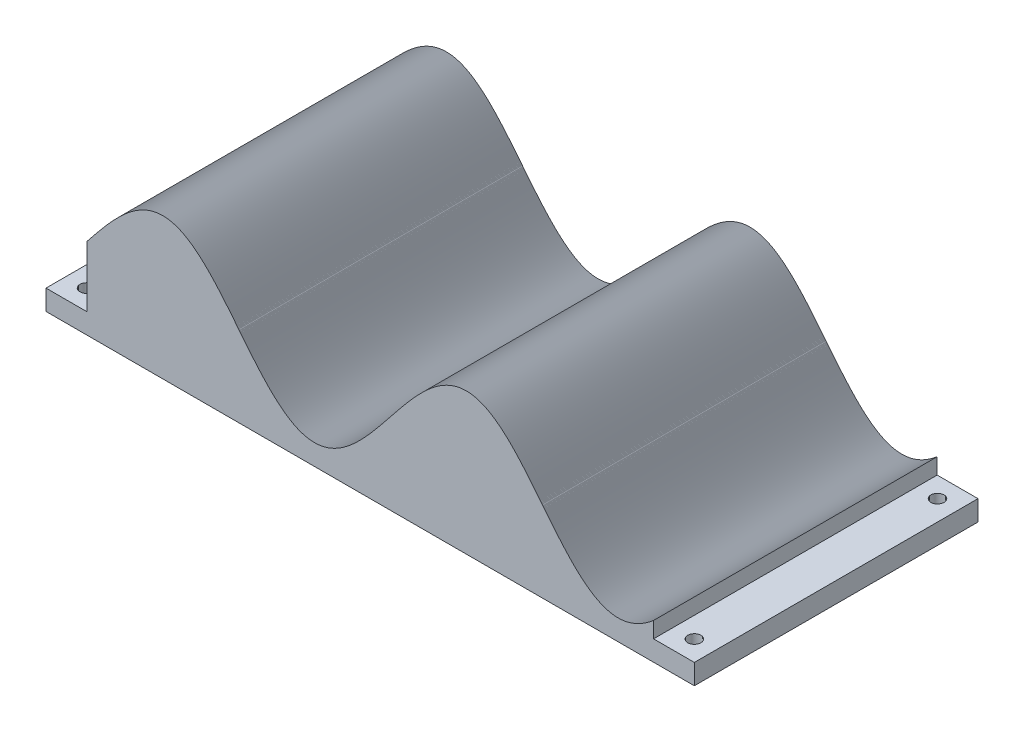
SolidWorks part; units mm, degrees
ref_plane "Front Plane" through (0, 0, 0) normal (0, 0, 1) x (1, 0, 0)
ref_plane "Top Plane" through (0, 0, 0) normal (0, 1, 0) x (1, 0, 0)
ref_plane "Right Plane" through (0, 0, 0) normal (1, 0, 0) x (0, 0, -1)
sketch "Model" plane through (0, 0, 0) normal (0, 0, 1) x (1, 0, 0)
  line L0 (0.1685, 30) -> (0.2684, 30.1247)
  line L1 (0.2684, 30.1247) -> (0.3683, 30.2495)
  line L2 (0.3683, 30.2495) -> (0.4682, 30.3743)
  line L3 (0.4682, 30.3743) -> (0.5681, 30.499)
  line L4 (0.5681, 30.499) -> (0.668, 30.6237)
  line L5 (0.668, 30.6237) -> (0.7679, 30.7485)
  line L6 (0.7679, 30.7485) -> (0.8678, 30.8732)
  line L7 (0.8678, 30.8732) -> (0.9676, 30.9979)
  line L8 (0.9676, 30.9979) -> (1.0675, 31.1226)
  line L9 (1.0675, 31.1226) -> (1.1674, 31.2472)
  line L10 (1.1674, 31.2472) -> (1.2673, 31.3719)
  line L11 (1.2673, 31.3719) -> (1.3672, 31.4965)
  line L12 (1.3672, 31.4965) -> (1.4671, 31.6211)
  line L13 (1.4671, 31.6211) -> (1.567, 31.7456)
  line L14 (1.567, 31.7456) -> (1.6669, 31.8702)
  line L15 (1.6669, 31.8702) -> (1.7668, 31.9947)
  line L16 (1.7668, 31.9947) -> (1.8667, 32.1191)
  line L17 (1.8667, 32.1191) -> (1.9665, 32.2435)
  line L18 (1.9665, 32.2435) -> (2.0664, 32.3679)
  line L19 (2.0664, 32.3679) -> (2.1663, 32.4923)
  line L20 (2.1663, 32.4923) -> (2.2662, 32.6166)
  line L21 (2.2662, 32.6166) -> (2.3661, 32.7408)
  line L22 (2.3661, 32.7408) -> (2.466, 32.865)
  line L23 (2.466, 32.865) -> (2.5659, 32.9892)
  line L24 (2.5659, 32.9892) -> (2.6658, 33.1133)
  line L25 (2.6658, 33.1133) -> (2.7657, 33.2374)
  line L26 (2.7657, 33.2374) -> (2.8656, 33.3613)
  line L27 (2.8656, 33.3613) -> (2.9654, 33.4853)
  line L28 (2.9654, 33.4853) -> (3.0653, 33.6091)
  line L29 (3.0653, 33.6091) -> (3.1652, 33.733)
  line L30 (3.1652, 33.733) -> (3.2651, 33.8567)
  line L31 (3.2651, 33.8567) -> (3.365, 33.9804)
  line L32 (3.365, 33.9804) -> (3.4649, 34.104)
  line L33 (3.4649, 34.104) -> (3.5648, 34.2275)
  line L34 (3.5648, 34.2275) -> (3.6647, 34.351)
  line L35 (3.6647, 34.351) -> (3.7646, 34.4743)
  line L36 (3.7646, 34.4743) -> (3.8645, 34.5976)
  line L37 (3.8645, 34.5976) -> (3.9643, 34.7209)
  line L38 (3.9643, 34.7209) -> (4.0642, 34.844)
  line L39 (4.0642, 34.844) -> (4.1641, 34.9671)
  line L40 (4.1641, 34.9671) -> (4.264, 35.09)
  line L41 (4.264, 35.09) -> (4.3639, 35.2129)
  line L42 (4.3639, 35.2129) -> (4.4638, 35.3357)
  line L43 (4.4638, 35.3357) -> (4.5637, 35.4584)
  line L44 (4.5637, 35.4584) -> (4.6636, 35.581)
  line L45 (4.6636, 35.581) -> (4.7635, 35.7035)
  line L46 (4.7635, 35.7035) -> (4.8634, 35.8259)
  line L47 (4.8634, 35.8259) -> (4.9633, 35.9482)
  line L48 (4.9633, 35.9482) -> (5.0631, 36.0704)
  line L49 (5.0631, 36.0704) -> (5.163, 36.1925)
  line L50 (5.163, 36.1925) -> (5.2629, 36.3145)
  line L51 (5.2629, 36.3145) -> (5.3628, 36.4363)
  line L52 (5.3628, 36.4363) -> (5.4627, 36.5581)
  line L53 (5.4627, 36.5581) -> (5.5626, 36.6797)
  line L54 (5.5626, 36.6797) -> (5.6625, 36.8013)
  line L55 (5.6625, 36.8013) -> (5.7624, 36.9227)
  line L56 (5.7624, 36.9227) -> (5.8623, 37.0439)
  line L57 (5.8623, 37.0439) -> (5.9622, 37.1651)
  line L58 (5.9622, 37.1651) -> (6.062, 37.2861)
  line L59 (6.062, 37.2861) -> (6.1619, 37.407)
  line L60 (6.1619, 37.407) -> (6.2618, 37.5278)
  line L61 (6.2618, 37.5278) -> (6.3617, 37.6485)
  line L62 (6.3617, 37.6485) -> (6.4616, 37.7689)
  line L63 (6.4616, 37.7689) -> (6.5615, 37.8893)
  line L64 (6.5615, 37.8893) -> (6.6614, 38.0095)
  line L65 (6.6614, 38.0095) -> (6.7613, 38.1296)
  line L66 (6.7613, 38.1296) -> (6.8612, 38.2496)
  line L67 (6.8612, 38.2496) -> (6.9611, 38.3694)
  line L68 (6.9611, 38.3694) -> (7.0609, 38.4891)
  line L69 (7.0609, 38.4891) -> (7.1608, 38.6086)
  line L70 (7.1608, 38.6086) -> (7.2607, 38.7279)
  line L71 (7.2607, 38.7279) -> (7.3606, 38.8471)
  line L72 (7.3606, 38.8471) -> (7.4605, 38.9662)
  line L73 (7.4605, 38.9662) -> (7.5604, 39.0851)
  line L74 (7.5604, 39.0851) -> (7.6603, 39.2038)
  line L75 (7.6603, 39.2038) -> (7.7602, 39.3224)
  line L76 (7.7602, 39.3224) -> (7.8601, 39.4408)
  line L77 (7.8601, 39.4408) -> (7.96, 39.559)
  line L78 (7.96, 39.559) -> (8.0598, 39.6771)
  line L79 (8.0598, 39.6771) -> (8.1597, 39.795)
  line L80 (8.1597, 39.795) -> (8.2596, 39.9128)
  line L81 (8.2596, 39.9128) -> (8.3595, 40.0303)
  line L82 (8.3595, 40.0303) -> (8.4594, 40.1477)
  line L83 (8.4594, 40.1477) -> (8.5593, 40.2649)
  line L84 (8.5593, 40.2649) -> (8.6592, 40.3819)
  line L85 (8.6592, 40.3819) -> (8.7591, 40.4988)
  line L86 (8.7591, 40.4988) -> (8.859, 40.6154)
  line L87 (8.859, 40.6154) -> (8.9589, 40.7319)
  line L88 (8.9589, 40.7319) -> (9.0587, 40.8482)
  line L89 (9.0587, 40.8482) -> (9.1586, 40.9643)
  line L90 (9.1586, 40.9643) -> (9.2585, 41.0802)
  line L91 (9.2585, 41.0802) -> (9.3584, 41.1959)
  line L92 (9.3584, 41.1959) -> (9.4583, 41.3114)
  line L93 (9.4583, 41.3114) -> (9.5582, 41.4267)
  line L94 (9.5582, 41.4267) -> (9.6581, 41.5418)
  line L95 (9.6581, 41.5418) -> (9.758, 41.6567)
  line L96 (9.758, 41.6567) -> (9.8579, 41.7715)
  line L97 (9.8579, 41.7715) -> (9.9578, 41.8859)
  line L98 (9.9578, 41.8859) -> (10.0576, 42.0002)
  line L99 (10.0576, 42.0002) -> (10.1575, 42.1143)
  line L100 (10.1575, 42.1143) -> (10.2574, 42.2282)
  line L101 (10.2574, 42.2282) -> (10.3573, 42.3419)
  line L102 (10.3573, 42.3419) -> (10.4572, 42.4553)
  line L103 (10.4572, 42.4553) -> (10.5571, 42.5685)
  line L104 (10.5571, 42.5685) -> (10.657, 42.6815)
  line L105 (10.657, 42.6815) -> (10.7569, 42.7943)
  line L106 (10.7569, 42.7943) -> (10.8568, 42.9068)
  line L107 (10.8568, 42.9068) -> (10.9567, 43.0191)
  line L108 (10.9567, 43.0191) -> (11.0565, 43.1312)
  line L109 (11.0565, 43.1312) -> (11.1564, 43.2431)
  line L110 (11.1564, 43.2431) -> (11.2563, 43.3548)
  line L111 (11.2563, 43.3548) -> (11.3562, 43.4661)
  line L112 (11.3562, 43.4661) -> (11.4561, 43.5773)
  line L113 (11.4561, 43.5773) -> (11.556, 43.6882)
  line L114 (11.556, 43.6882) -> (11.6559, 43.7989)
  line L115 (11.6559, 43.7989) -> (11.7558, 43.9093)
  line L116 (11.7558, 43.9093) -> (11.8557, 44.0195)
  line L117 (11.8557, 44.0195) -> (11.9556, 44.1295)
  line L118 (11.9556, 44.1295) -> (12.0554, 44.2392)
  line L119 (12.0554, 44.2392) -> (12.1553, 44.3487)
  line L120 (12.1553, 44.3487) -> (12.2552, 44.4578)
  line L121 (12.2552, 44.4578) -> (12.3551, 44.5668)
  line L122 (12.3551, 44.5668) -> (12.455, 44.6755)
  line L123 (12.455, 44.6755) -> (12.5549, 44.7839)
  line L124 (12.5549, 44.7839) -> (12.6548, 44.8921)
  line L125 (12.6548, 44.8921) -> (12.7547, 45)
  line L126 (12.7547, 45) -> (12.8546, 45.1077)
  line L127 (12.8546, 45.1077) -> (12.9545, 45.2151)
  line L128 (12.9545, 45.2151) -> (13.0543, 45.3222)
  line L129 (13.0543, 45.3222) -> (13.1542, 45.429)
  line L130 (13.1542, 45.429) -> (13.2541, 45.5356)
  line L131 (13.2541, 45.5356) -> (13.354, 45.6419)
  line L132 (13.354, 45.6419) -> (13.4539, 45.7479)
  line L133 (13.4539, 45.7479) -> (13.5538, 45.8537)
  line L134 (13.5538, 45.8537) -> (13.6537, 45.9592)
  line L135 (13.6537, 45.9592) -> (13.7536, 46.0644)
  line L136 (13.7536, 46.0644) -> (13.8535, 46.1693)
  line L137 (13.8535, 46.1693) -> (13.9534, 46.2739)
  line L138 (13.9534, 46.2739) -> (14.0533, 46.3783)
  line L139 (14.0533, 46.3783) -> (14.1531, 46.4823)
  line L140 (14.1531, 46.4823) -> (14.253, 46.5861)
  line L141 (14.253, 46.5861) -> (14.3529, 46.6896)
  line L142 (14.3529, 46.6896) -> (14.4528, 46.7928)
  line L143 (14.4528, 46.7928) -> (14.5527, 46.8957)
  line L144 (14.5527, 46.8957) -> (14.6526, 46.9982)
  line L145 (14.6526, 46.9982) -> (14.7525, 47.1005)
  line L146 (14.7525, 47.1005) -> (14.8524, 47.2025)
  line L147 (14.8524, 47.2025) -> (14.9523, 47.3042)
  line L148 (14.9523, 47.3042) -> (15.0522, 47.4056)
  line L149 (15.0522, 47.4056) -> (15.152, 47.5067)
  line L150 (15.152, 47.5067) -> (15.2519, 47.6075)
  line L151 (15.2519, 47.6075) -> (15.3518, 47.708)
  line L152 (15.3518, 47.708) -> (15.4517, 47.8081)
  line L153 (15.4517, 47.8081) -> (15.5516, 47.908)
  line L154 (15.5516, 47.908) -> (15.6515, 48.0075)
  line L155 (15.6515, 48.0075) -> (15.7514, 48.1067)
  line L156 (15.7514, 48.1067) -> (15.8513, 48.2056)
  line L157 (15.8513, 48.2056) -> (15.9512, 48.3042)
  line L158 (15.9512, 48.3042) -> (16.0511, 48.4024)
  line L159 (16.0511, 48.4024) -> (16.1509, 48.5004)
  line L160 (16.1509, 48.5004) -> (16.2508, 48.598)
  line L161 (16.2508, 48.598) -> (16.3507, 48.6953)
  line L162 (16.3507, 48.6953) -> (16.4506, 48.7922)
  line L163 (16.4506, 48.7922) -> (16.5505, 48.8889)
  line L164 (16.5505, 48.8889) -> (16.6504, 48.9852)
  line L165 (16.6504, 48.9852) -> (16.7503, 49.0811)
  line L166 (16.7503, 49.0811) -> (16.8502, 49.1768)
  line L167 (16.8502, 49.1768) -> (16.9501, 49.272)
  line L168 (16.9501, 49.272) -> (17.05, 49.367)
  line L169 (17.05, 49.367) -> (17.1498, 49.4616)
  line L170 (17.1498, 49.4616) -> (17.2497, 49.5559)
  line L171 (17.2497, 49.5559) -> (17.3496, 49.6498)
  line L172 (17.3496, 49.6498) -> (17.4495, 49.7434)
  line L173 (17.4495, 49.7434) -> (17.5494, 49.8366)
  line L174 (17.5494, 49.8366) -> (17.6493, 49.9295)
  line L175 (17.6493, 49.9295) -> (17.7492, 50.022)
  line L176 (17.7492, 50.022) -> (17.8491, 50.1143)
  line L177 (17.8491, 50.1143) -> (17.949, 50.2061)
  line L178 (17.949, 50.2061) -> (18.0489, 50.2976)
  line L179 (18.0489, 50.2976) -> (18.1487, 50.3887)
  line L180 (18.1487, 50.3887) -> (18.2486, 50.4794)
  line L181 (18.2486, 50.4794) -> (18.3485, 50.5699)
  line L182 (18.3485, 50.5699) -> (18.4484, 50.6599)
  line L183 (18.4484, 50.6599) -> (18.5483, 50.7496)
  line L184 (18.5483, 50.7496) -> (18.6482, 50.8389)
  line L185 (18.6482, 50.8389) -> (18.7481, 50.9279)
  line L186 (18.7481, 50.9279) -> (18.848, 51.0164)
  line L187 (18.848, 51.0164) -> (18.9479, 51.1047)
  line L188 (18.9479, 51.1047) -> (19.0478, 51.1925)
  line L189 (19.0478, 51.1925) -> (19.1476, 51.28)
  line L190 (19.1476, 51.28) -> (19.2475, 51.3671)
  line L191 (19.2475, 51.3671) -> (19.3474, 51.4538)
  line L192 (19.3474, 51.4538) -> (19.4473, 51.5402)
  line L193 (19.4473, 51.5402) -> (19.5472, 51.6262)
  line L194 (19.5472, 51.6262) -> (19.6471, 51.7118)
  line L195 (19.6471, 51.7118) -> (19.747, 51.797)
  line L196 (19.747, 51.797) -> (19.8469, 51.8818)
  line L197 (19.8469, 51.8818) -> (19.9468, 51.9662)
  line L198 (19.9468, 51.9662) -> (20.0467, 52.0503)
  line L199 (20.0467, 52.0503) -> (20.1465, 52.134)
  line L200 (20.1465, 52.134) -> (20.2464, 52.2173)
  line L201 (20.2464, 52.2173) -> (20.3463, 52.3001)
  line L202 (20.3463, 52.3001) -> (20.4462, 52.3827)
  line L203 (20.4462, 52.3827) -> (20.5461, 52.4648)
  line L204 (20.5461, 52.4648) -> (20.646, 52.5465)
  line L205 (20.646, 52.5465) -> (20.7459, 52.6278)
  line L206 (20.7459, 52.6278) -> (20.8458, 52.7087)
  line L207 (20.8458, 52.7087) -> (20.9457, 52.7893)
  line L208 (20.9457, 52.7893) -> (21.0456, 52.8694)
  line L209 (21.0456, 52.8694) -> (21.1454, 52.9491)
  line L210 (21.1454, 52.9491) -> (21.2453, 53.0284)
  line L211 (21.2453, 53.0284) -> (21.3452, 53.1074)
  line L212 (21.3452, 53.1074) -> (21.4451, 53.1859)
  line L213 (21.4451, 53.1859) -> (21.545, 53.264)
  line L214 (21.545, 53.264) -> (21.6449, 53.3417)
  line L215 (21.6449, 53.3417) -> (21.7448, 53.419)
  line L216 (21.7448, 53.419) -> (21.8447, 53.4958)
  line L217 (21.8447, 53.4958) -> (21.9446, 53.5723)
  line L218 (21.9446, 53.5723) -> (22.0445, 53.6484)
  line L219 (22.0445, 53.6484) -> (22.1443, 53.724)
  line L220 (22.1443, 53.724) -> (22.2442, 53.7992)
  line L221 (22.2442, 53.7992) -> (22.3441, 53.874)
  line L222 (22.3441, 53.874) -> (22.444, 53.9484)
  line L223 (22.444, 53.9484) -> (22.5439, 54.0224)
  line L224 (22.5439, 54.0224) -> (22.6438, 54.0959)
  line L225 (22.6438, 54.0959) -> (22.7437, 54.169)
  line L226 (22.7437, 54.169) -> (22.8436, 54.2418)
  line L227 (22.8436, 54.2418) -> (22.9435, 54.314)
  line L228 (22.9435, 54.314) -> (23.0434, 54.3858)
  line L229 (23.0434, 54.3858) -> (23.1432, 54.4573)
  line L230 (23.1432, 54.4573) -> (23.2431, 54.5283)
  line L231 (23.2431, 54.5283) -> (23.343, 54.5988)
  line L232 (23.343, 54.5988) -> (23.4429, 54.6689)
  line L233 (23.4429, 54.6689) -> (23.5428, 54.7386)
  line L234 (23.5428, 54.7386) -> (23.6427, 54.8079)
  line L235 (23.6427, 54.8079) -> (23.7426, 54.8767)
  line L236 (23.7426, 54.8767) -> (23.8425, 54.9451)
  line L237 (23.8425, 54.9451) -> (23.9424, 55.013)
  line L238 (23.9424, 55.013) -> (24.0423, 55.0806)
  line L239 (24.0423, 55.0806) -> (24.1422, 55.1476)
  line L240 (24.1422, 55.1476) -> (24.242, 55.2142)
  line L241 (24.242, 55.2142) -> (24.3419, 55.2804)
  line L242 (24.3419, 55.2804) -> (24.4418, 55.3462)
  line L243 (24.4418, 55.3462) -> (24.5417, 55.4115)
  line L244 (24.5417, 55.4115) -> (24.6416, 55.4763)
  line L245 (24.6416, 55.4763) -> (24.7415, 55.5407)
  line L246 (24.7415, 55.5407) -> (24.8414, 55.6047)
  line L247 (24.8414, 55.6047) -> (24.9413, 55.6682)
  line L248 (24.9413, 55.6682) -> (25.0412, 55.7313)
  line L249 (25.0412, 55.7313) -> (25.1411, 55.7939)
  line L250 (25.1411, 55.7939) -> (25.2409, 55.856)
  line L251 (25.2409, 55.856) -> (25.3408, 55.9177)
  line L252 (25.3408, 55.9177) -> (25.4407, 55.979)
  line L253 (25.4407, 55.979) -> (25.5406, 56.0397)
  line L254 (25.5406, 56.0397) -> (25.6405, 56.1001)
  line L255 (25.6405, 56.1001) -> (25.7404, 56.16)
  line L256 (25.7404, 56.16) -> (25.8403, 56.2194)
  line L257 (25.8403, 56.2194) -> (25.9402, 56.2783)
  line L258 (25.9402, 56.2783) -> (26.0401, 56.3368)
  line L259 (26.0401, 56.3368) -> (26.14, 56.3949)
  line L260 (26.14, 56.3949) -> (26.2398, 56.4524)
  line L261 (26.2398, 56.4524) -> (26.3397, 56.5095)
  line L262 (26.3397, 56.5095) -> (26.4396, 56.5662)
  line L263 (26.4396, 56.5662) -> (26.5395, 56.6224)
  line L264 (26.5395, 56.6224) -> (26.6394, 56.678)
  line L265 (26.6394, 56.678) -> (26.7393, 56.7333)
  line L266 (26.7393, 56.7333) -> (26.8392, 56.788)
  line L267 (26.8392, 56.788) -> (26.9391, 56.8424)
  line L268 (26.9391, 56.8424) -> (27.039, 56.8962)
  line L269 (27.039, 56.8962) -> (27.1389, 56.9495)
  line L270 (27.1389, 56.9495) -> (27.2387, 57.0024)
  line L271 (27.2387, 57.0024) -> (27.3386, 57.0548)
  line L272 (27.3386, 57.0548) -> (27.4385, 57.1068)
  line L273 (27.4385, 57.1068) -> (27.5384, 57.1582)
  line L274 (27.5384, 57.1582) -> (27.6383, 57.2092)
  line L275 (27.6383, 57.2092) -> (27.7382, 57.2597)
  line L276 (27.7382, 57.2597) -> (27.8381, 57.3098)
  line L277 (27.8381, 57.3098) -> (27.938, 57.3593)
  line L278 (27.938, 57.3593) -> (28.0379, 57.4084)
  line L279 (28.0379, 57.4084) -> (28.1378, 57.457)
  line L280 (28.1378, 57.457) -> (28.2376, 57.5051)
  line L281 (28.2376, 57.5051) -> (28.3375, 57.5527)
  line L282 (28.3375, 57.5527) -> (28.4374, 57.5998)
  line L283 (28.4374, 57.5998) -> (28.5373, 57.6465)
  line L284 (28.5373, 57.6465) -> (28.6372, 57.6927)
  line L285 (28.6372, 57.6927) -> (28.7371, 57.7383)
  line L286 (28.7371, 57.7383) -> (28.837, 57.7835)
  line L287 (28.837, 57.7835) -> (28.9369, 57.8282)
  line L288 (28.9369, 57.8282) -> (29.0368, 57.8725)
  line L289 (29.0368, 57.8725) -> (29.1367, 57.9162)
  line L290 (29.1367, 57.9162) -> (29.2366, 57.9594)
  line L291 (29.2366, 57.9594) -> (29.3364, 58.0022)
  line L292 (29.3364, 58.0022) -> (29.4363, 58.0444)
  line L293 (29.4363, 58.0444) -> (29.5362, 58.0862)
  line L294 (29.5362, 58.0862) -> (29.6361, 58.1275)
  line L295 (29.6361, 58.1275) -> (29.736, 58.1683)
  line L296 (29.736, 58.1683) -> (29.8359, 58.2086)
  line L297 (29.8359, 58.2086) -> (29.9358, 58.2484)
  line L298 (29.9358, 58.2484) -> (30.0357, 58.2877)
  line L299 (30.0357, 58.2877) -> (30.1356, 58.3265)
  line L300 (30.1356, 58.3265) -> (30.2354, 58.3648)
  line L301 (30.2354, 58.3648) -> (30.3353, 58.4026)
  line L302 (30.3353, 58.4026) -> (30.4352, 58.4399)
  line L303 (30.4352, 58.4399) -> (30.5351, 58.4767)
  line L304 (30.5351, 58.4767) -> (30.635, 58.513)
  line L305 (30.635, 58.513) -> (30.7349, 58.5488)
  line L306 (30.7349, 58.5488) -> (30.8348, 58.5841)
  line L307 (30.8348, 58.5841) -> (30.9347, 58.6189)
  line L308 (30.9347, 58.6189) -> (31.0346, 58.6532)
  line L309 (31.0346, 58.6532) -> (31.1345, 58.687)
  line L310 (31.1345, 58.687) -> (31.2343, 58.7203)
  line L311 (31.2343, 58.7203) -> (31.3342, 58.7531)
  line L312 (31.3342, 58.7531) -> (31.4341, 58.7854)
  line L313 (31.4341, 58.7854) -> (31.534, 58.8172)
  line L314 (31.534, 58.8172) -> (31.6339, 58.8485)
  line L315 (31.6339, 58.8485) -> (31.7338, 58.8792)
  line L316 (31.7338, 58.8792) -> (31.8337, 58.9095)
  line L317 (31.8337, 58.9095) -> (31.9336, 58.9393)
  line L318 (31.9336, 58.9393) -> (32.0335, 58.9685)
  line L319 (32.0335, 58.9685) -> (32.1334, 58.9973)
  line L320 (32.1334, 58.9973) -> (32.2333, 59.0255)
  line L321 (32.2333, 59.0255) -> (32.3331, 59.0532)
  line L322 (32.3331, 59.0532) -> (32.433, 59.0804)
  line L323 (32.433, 59.0804) -> (32.5329, 59.1071)
  line L324 (32.5329, 59.1071) -> (32.6328, 59.1333)
  line L325 (32.6328, 59.1333) -> (32.7327, 59.159)
  line L326 (32.7327, 59.159) -> (32.8326, 59.1842)
  line L327 (32.8326, 59.1842) -> (32.9325, 59.2089)
  line L328 (32.9325, 59.2089) -> (33.0324, 59.233)
  line L329 (33.0324, 59.233) -> (33.1323, 59.2566)
  line L330 (33.1323, 59.2566) -> (33.2322, 59.2797)
  line L331 (33.2322, 59.2797) -> (33.332, 59.3024)
  line L332 (33.332, 59.3024) -> (33.4319, 59.3245)
  line L333 (33.4319, 59.3245) -> (33.5318, 59.346)
  line L334 (33.5318, 59.346) -> (33.6317, 59.3671)
  line L335 (33.6317, 59.3671) -> (33.7316, 59.3877)
  line L336 (33.7316, 59.3877) -> (33.8315, 59.4077)
  line L337 (33.8315, 59.4077) -> (33.9314, 59.4272)
  line L338 (33.9314, 59.4272) -> (34.0313, 59.4462)
  line L339 (34.0313, 59.4462) -> (34.1312, 59.4647)
  line L340 (34.1312, 59.4647) -> (34.2311, 59.4826)
  line L341 (34.2311, 59.4826) -> (34.3309, 59.5001)
  line L342 (34.3309, 59.5001) -> (34.4308, 59.517)
  line L343 (34.4308, 59.517) -> (34.5307, 59.5334)
  line L344 (34.5307, 59.5334) -> (34.6306, 59.5493)
  line L345 (34.6306, 59.5493) -> (34.7305, 59.5647)
  line L346 (34.7305, 59.5647) -> (34.8304, 59.5796)
  line L347 (34.8304, 59.5796) -> (34.9303, 59.5939)
  line L348 (34.9303, 59.5939) -> (35.0302, 59.6077)
  line L349 (35.0302, 59.6077) -> (35.1301, 59.621)
  line L350 (35.1301, 59.621) -> (35.2299, 59.6338)
  line L351 (35.2299, 59.6338) -> (35.3298, 59.6461)
  line L352 (35.3298, 59.6461) -> (35.4297, 59.6578)
  line L353 (35.4297, 59.6578) -> (35.5296, 59.669)
  line L354 (35.5296, 59.669) -> (35.6295, 59.6798)
  line L355 (35.6295, 59.6798) -> (35.7294, 59.6899)
  line L356 (35.7294, 59.6899) -> (35.8293, 59.6996)
  line L357 (35.8293, 59.6996) -> (35.9292, 59.7087)
  line L358 (35.9292, 59.7087) -> (36.0291, 59.7173)
  line L359 (36.0291, 59.7173) -> (36.129, 59.7254)
  line L360 (36.129, 59.7254) -> (36.2289, 59.733)
  line L361 (36.2289, 59.733) -> (36.3287, 59.7401)
  line L362 (36.3287, 59.7401) -> (36.4286, 59.7466)
  line L363 (36.4286, 59.7466) -> (36.5285, 59.7526)
  line L364 (36.5285, 59.7526) -> (36.6284, 59.7581)
  line L365 (36.6284, 59.7581) -> (36.7283, 59.763)
  line L366 (36.7283, 59.763) -> (36.8282, 59.7675)
  line L367 (36.8282, 59.7675) -> (36.9281, 59.7714)
  line L368 (36.9281, 59.7714) -> (37.028, 59.7748)
  line L369 (37.028, 59.7748) -> (37.1279, 59.7777)
  line L370 (37.1279, 59.7777) -> (37.2278, 59.78)
  line L371 (37.2278, 59.78) -> (37.3276, 59.7819)
  line L372 (37.3276, 59.7819) -> (37.4275, 59.7832)
  line L373 (37.4275, 59.7832) -> (37.5274, 59.7839)
  line L374 (37.5274, 59.7839) -> (37.6273, 59.7841)
  line L375 (37.6273, 59.7841) -> (37.7272, 59.7839)
  line L376 (37.7272, 59.7839) -> (37.8271, 59.7832)
  line L377 (37.8271, 59.7832) -> (37.927, 59.7819)
  line L378 (37.927, 59.7819) -> (38.0269, 59.78)
  line L379 (38.0269, 59.78) -> (38.1268, 59.7777)
  line L380 (38.1268, 59.7777) -> (38.2267, 59.7748)
  line L381 (38.2267, 59.7748) -> (38.3265, 59.7714)
  line L382 (38.3265, 59.7714) -> (38.4264, 59.7675)
  line L383 (38.4264, 59.7675) -> (38.5263, 59.763)
  line L384 (38.5263, 59.763) -> (38.6262, 59.7581)
  line L385 (38.6262, 59.7581) -> (38.7261, 59.7526)
  line L386 (38.7261, 59.7526) -> (38.826, 59.7466)
  line L387 (38.826, 59.7466) -> (38.9259, 59.7401)
  line L388 (38.9259, 59.7401) -> (39.0258, 59.733)
  line L389 (39.0258, 59.733) -> (39.1257, 59.7254)
  line L390 (39.1257, 59.7254) -> (39.2256, 59.7173)
  line L391 (39.2256, 59.7173) -> (39.3255, 59.7087)
  line L392 (39.3255, 59.7087) -> (39.4253, 59.6996)
  line L393 (39.4253, 59.6996) -> (39.5252, 59.6899)
  line L394 (39.5252, 59.6899) -> (39.6251, 59.6798)
  line L395 (39.6251, 59.6798) -> (39.725, 59.669)
  line L396 (39.725, 59.669) -> (39.8249, 59.6578)
  line L397 (39.8249, 59.6578) -> (39.9248, 59.6461)
  line L398 (39.9248, 59.6461) -> (40.0247, 59.6338)
  line L399 (40.0247, 59.6338) -> (40.1246, 59.621)
  line L400 (40.1246, 59.621) -> (40.2245, 59.6077)
  line L401 (40.2245, 59.6077) -> (40.3243, 59.5939)
  line L402 (40.3243, 59.5939) -> (40.4242, 59.5796)
  line L403 (40.4242, 59.5796) -> (40.5241, 59.5647)
  line L404 (40.5241, 59.5647) -> (40.624, 59.5493)
  line L405 (40.624, 59.5493) -> (40.7239, 59.5334)
  line L406 (40.7239, 59.5334) -> (40.8238, 59.517)
  line L407 (40.8238, 59.517) -> (40.9237, 59.5001)
  line L408 (40.9237, 59.5001) -> (41.0236, 59.4826)
  line L409 (41.0236, 59.4826) -> (41.1235, 59.4647)
  line L410 (41.1235, 59.4647) -> (41.2234, 59.4462)
  line L411 (41.2234, 59.4462) -> (41.3232, 59.4272)
  line L412 (41.3232, 59.4272) -> (41.4231, 59.4077)
  line L413 (41.4231, 59.4077) -> (41.523, 59.3877)
  line L414 (41.523, 59.3877) -> (41.6229, 59.3671)
  line L415 (41.6229, 59.3671) -> (41.7228, 59.346)
  line L416 (41.7228, 59.346) -> (41.8227, 59.3245)
  line L417 (41.8227, 59.3245) -> (41.9226, 59.3024)
  line L418 (41.9226, 59.3024) -> (42.0225, 59.2797)
  line L419 (42.0225, 59.2797) -> (42.1224, 59.2566)
  line L420 (42.1224, 59.2566) -> (42.2223, 59.233)
  line L421 (42.2223, 59.233) -> (42.3221, 59.2089)
  line L422 (42.3221, 59.2089) -> (42.422, 59.1842)
  line L423 (42.422, 59.1842) -> (42.5219, 59.159)
  line L424 (42.5219, 59.159) -> (42.6218, 59.1333)
  line L425 (42.6218, 59.1333) -> (42.7217, 59.1071)
  line L426 (42.7217, 59.1071) -> (42.8216, 59.0804)
  line L427 (42.8216, 59.0804) -> (42.9215, 59.0532)
  line L428 (42.9215, 59.0532) -> (43.0214, 59.0255)
  line L429 (43.0214, 59.0255) -> (43.1213, 58.9973)
  line L430 (43.1213, 58.9973) -> (43.2212, 58.9685)
  line L431 (43.2212, 58.9685) -> (43.3211, 58.9393)
  line L432 (43.3211, 58.9393) -> (43.4209, 58.9095)
  line L433 (43.4209, 58.9095) -> (43.5208, 58.8792)
  line L434 (43.5208, 58.8792) -> (43.6207, 58.8485)
  line L435 (43.6207, 58.8485) -> (43.7206, 58.8172)
  line L436 (43.7206, 58.8172) -> (43.8205, 58.7854)
  line L437 (43.8205, 58.7854) -> (43.9204, 58.7531)
  line L438 (43.9204, 58.7531) -> (44.0203, 58.7203)
  line L439 (44.0203, 58.7203) -> (44.1202, 58.687)
  line L440 (44.1202, 58.687) -> (44.2201, 58.6532)
  line L441 (44.2201, 58.6532) -> (44.32, 58.6189)
  line L442 (44.32, 58.6189) -> (44.4198, 58.5841)
  line L443 (44.4198, 58.5841) -> (44.5197, 58.5488)
  line L444 (44.5197, 58.5488) -> (44.6196, 58.513)
  line L445 (44.6196, 58.513) -> (44.7195, 58.4767)
  line L446 (44.7195, 58.4767) -> (44.8194, 58.4399)
  line L447 (44.8194, 58.4399) -> (44.9193, 58.4026)
  line L448 (44.9193, 58.4026) -> (45.0192, 58.3648)
  line L449 (45.0192, 58.3648) -> (45.1191, 58.3265)
  line L450 (45.1191, 58.3265) -> (45.219, 58.2877)
  line L451 (45.219, 58.2877) -> (45.3189, 58.2484)
  line L452 (45.3189, 58.2484) -> (45.4187, 58.2086)
  line L453 (45.4187, 58.2086) -> (45.5186, 58.1683)
  line L454 (45.5186, 58.1683) -> (45.6185, 58.1275)
  line L455 (45.6185, 58.1275) -> (45.7184, 58.0862)
  line L456 (45.7184, 58.0862) -> (45.8183, 58.0444)
  line L457 (45.8183, 58.0444) -> (45.9182, 58.0022)
  line L458 (45.9182, 58.0022) -> (46.0181, 57.9594)
  line L459 (46.0181, 57.9594) -> (46.118, 57.9162)
  line L460 (46.118, 57.9162) -> (46.2179, 57.8725)
  line L461 (46.2179, 57.8725) -> (46.3178, 57.8282)
  line L462 (46.3178, 57.8282) -> (46.4176, 57.7835)
  line L463 (46.4176, 57.7835) -> (46.5175, 57.7383)
  line L464 (46.5175, 57.7383) -> (46.6174, 57.6927)
  line L465 (46.6174, 57.6927) -> (46.7173, 57.6465)
  line L466 (46.7173, 57.6465) -> (46.8172, 57.5998)
  line L467 (46.8172, 57.5998) -> (46.9171, 57.5527)
  line L468 (46.9171, 57.5527) -> (47.017, 57.5051)
  line L469 (47.017, 57.5051) -> (47.1169, 57.457)
  line L470 (47.1169, 57.457) -> (47.2168, 57.4084)
  line L471 (47.2168, 57.4084) -> (47.3167, 57.3593)
  line L472 (47.3167, 57.3593) -> (47.4165, 57.3098)
  line L473 (47.4165, 57.3098) -> (47.5164, 57.2597)
  line L474 (47.5164, 57.2597) -> (47.6163, 57.2092)
  line L475 (47.6163, 57.2092) -> (47.7162, 57.1582)
  line L476 (47.7162, 57.1582) -> (47.8161, 57.1068)
  line L477 (47.8161, 57.1068) -> (47.916, 57.0548)
  line L478 (47.916, 57.0548) -> (48.0159, 57.0024)
  line L479 (48.0159, 57.0024) -> (48.1158, 56.9495)
  line L480 (48.1158, 56.9495) -> (48.2157, 56.8962)
  line L481 (48.2157, 56.8962) -> (48.3156, 56.8424)
  line L482 (48.3156, 56.8424) -> (48.4154, 56.788)
  line L483 (48.4154, 56.788) -> (48.5153, 56.7333)
  line L484 (48.5153, 56.7333) -> (48.6152, 56.678)
  line L485 (48.6152, 56.678) -> (48.7151, 56.6224)
  line L486 (48.7151, 56.6224) -> (48.815, 56.5662)
  line L487 (48.815, 56.5662) -> (48.9149, 56.5095)
  line L488 (48.9149, 56.5095) -> (49.0148, 56.4524)
  line L489 (49.0148, 56.4524) -> (49.1147, 56.3949)
  line L490 (49.1147, 56.3949) -> (49.2146, 56.3368)
  line L491 (49.2146, 56.3368) -> (49.3145, 56.2783)
  line L492 (49.3145, 56.2783) -> (49.4143, 56.2194)
  line L493 (49.4143, 56.2194) -> (49.5142, 56.16)
  line L494 (49.5142, 56.16) -> (49.6141, 56.1001)
  line L495 (49.6141, 56.1001) -> (49.714, 56.0397)
  line L496 (49.714, 56.0397) -> (49.8139, 55.979)
  line L497 (49.8139, 55.979) -> (49.9138, 55.9177)
  line L498 (49.9138, 55.9177) -> (50.0137, 55.856)
  line L499 (50.0137, 55.856) -> (50.1136, 55.7939)
  line L500 (50.1136, 55.7939) -> (50.2135, 55.7313)
  line L501 (50.2135, 55.7313) -> (50.3134, 55.6682)
  line L502 (50.3134, 55.6682) -> (50.4133, 55.6047)
  line L503 (50.4133, 55.6047) -> (50.5131, 55.5407)
  line L504 (50.5131, 55.5407) -> (50.613, 55.4763)
  line L505 (50.613, 55.4763) -> (50.7129, 55.4115)
  line L506 (50.7129, 55.4115) -> (50.8128, 55.3462)
  line L507 (50.8128, 55.3462) -> (50.9127, 55.2804)
  line L508 (50.9127, 55.2804) -> (51.0126, 55.2142)
  line L509 (51.0126, 55.2142) -> (51.1125, 55.1476)
  line L510 (51.1125, 55.1476) -> (51.2124, 55.0806)
  line L511 (51.2124, 55.0806) -> (51.3123, 55.013)
  line L512 (51.3123, 55.013) -> (51.4122, 54.9451)
  line L513 (51.4122, 54.9451) -> (51.512, 54.8767)
  line L514 (51.512, 54.8767) -> (51.6119, 54.8079)
  line L515 (51.6119, 54.8079) -> (51.7118, 54.7386)
  line L516 (51.7118, 54.7386) -> (51.8117, 54.6689)
  line L517 (51.8117, 54.6689) -> (51.9116, 54.5988)
  line L518 (51.9116, 54.5988) -> (52.0115, 54.5283)
  line L519 (52.0115, 54.5283) -> (52.1114, 54.4573)
  line L520 (52.1114, 54.4573) -> (52.2113, 54.3858)
  line L521 (52.2113, 54.3858) -> (52.3112, 54.314)
  line L522 (52.3112, 54.314) -> (52.4111, 54.2418)
  line L523 (52.4111, 54.2418) -> (52.5109, 54.169)
  line L524 (52.5109, 54.169) -> (52.6108, 54.0959)
  line L525 (52.6108, 54.0959) -> (52.7107, 54.0224)
  line L526 (52.7107, 54.0224) -> (52.8106, 53.9484)
  line L527 (52.8106, 53.9484) -> (52.9105, 53.874)
  line L528 (52.9105, 53.874) -> (53.0104, 53.7992)
  line L529 (53.0104, 53.7992) -> (53.1103, 53.724)
  line L530 (53.1103, 53.724) -> (53.2102, 53.6484)
  line L531 (53.2102, 53.6484) -> (53.3101, 53.5723)
  line L532 (53.3101, 53.5723) -> (53.41, 53.4958)
  line L533 (53.41, 53.4958) -> (53.5098, 53.419)
  line L534 (53.5098, 53.419) -> (53.6097, 53.3417)
  line L535 (53.6097, 53.3417) -> (53.7096, 53.264)
  line L536 (53.7096, 53.264) -> (53.8095, 53.1859)
  line L537 (53.8095, 53.1859) -> (53.9094, 53.1074)
  line L538 (53.9094, 53.1074) -> (54.0093, 53.0284)
  line L539 (54.0093, 53.0284) -> (54.1092, 52.9491)
  line L540 (54.1092, 52.9491) -> (54.2091, 52.8694)
  line L541 (54.2091, 52.8694) -> (54.309, 52.7893)
  line L542 (54.309, 52.7893) -> (54.4089, 52.7087)
  line L543 (54.4089, 52.7087) -> (54.5087, 52.6278)
  line L544 (54.5087, 52.6278) -> (54.6086, 52.5465)
  line L545 (54.6086, 52.5465) -> (54.7085, 52.4648)
  line L546 (54.7085, 52.4648) -> (54.8084, 52.3827)
  line L547 (54.8084, 52.3827) -> (54.9083, 52.3001)
  line L548 (54.9083, 52.3001) -> (55.0082, 52.2173)
  line L549 (55.0082, 52.2173) -> (55.1081, 52.134)
  line L550 (55.1081, 52.134) -> (55.208, 52.0503)
  line L551 (55.208, 52.0503) -> (55.3079, 51.9662)
  line L552 (55.3079, 51.9662) -> (55.4078, 51.8818)
  line L553 (55.4078, 51.8818) -> (55.5076, 51.797)
  line L554 (55.5076, 51.797) -> (55.6075, 51.7118)
  line L555 (55.6075, 51.7118) -> (55.7074, 51.6262)
  line L556 (55.7074, 51.6262) -> (55.8073, 51.5402)
  line L557 (55.8073, 51.5402) -> (55.9072, 51.4538)
  line L558 (55.9072, 51.4538) -> (56.0071, 51.3671)
  line L559 (56.0071, 51.3671) -> (56.107, 51.28)
  line L560 (56.107, 51.28) -> (56.2069, 51.1925)
  line L561 (56.2069, 51.1925) -> (56.3068, 51.1047)
  line L562 (56.3068, 51.1047) -> (56.4067, 51.0164)
  line L563 (56.4067, 51.0164) -> (56.5065, 50.9279)
  line L564 (56.5065, 50.9279) -> (56.6064, 50.8389)
  line L565 (56.6064, 50.8389) -> (56.7063, 50.7496)
  line L566 (56.7063, 50.7496) -> (56.8062, 50.6599)
  line L567 (56.8062, 50.6599) -> (56.9061, 50.5699)
  line L568 (56.9061, 50.5699) -> (57.006, 50.4794)
  line L569 (57.006, 50.4794) -> (57.1059, 50.3887)
  line L570 (57.1059, 50.3887) -> (57.2058, 50.2976)
  line L571 (57.2058, 50.2976) -> (57.3057, 50.2061)
  line L572 (57.3057, 50.2061) -> (57.4056, 50.1143)
  line L573 (57.4056, 50.1143) -> (57.5054, 50.022)
  line L574 (57.5054, 50.022) -> (57.6053, 49.9295)
  line L575 (57.6053, 49.9295) -> (57.7052, 49.8366)
  line L576 (57.7052, 49.8366) -> (57.8051, 49.7434)
  line L577 (57.8051, 49.7434) -> (57.905, 49.6498)
  line L578 (57.905, 49.6498) -> (58.0049, 49.5559)
  line L579 (58.0049, 49.5559) -> (58.1048, 49.4616)
  line L580 (58.1048, 49.4616) -> (58.2047, 49.367)
  line L581 (58.2047, 49.367) -> (58.3046, 49.272)
  line L582 (58.3046, 49.272) -> (58.4045, 49.1768)
  line L583 (58.4045, 49.1768) -> (58.5043, 49.0811)
  line L584 (58.5043, 49.0811) -> (58.6042, 48.9852)
  line L585 (58.6042, 48.9852) -> (58.7041, 48.8889)
  line L586 (58.7041, 48.8889) -> (58.804, 48.7922)
  line L587 (58.804, 48.7922) -> (58.9039, 48.6953)
  line L588 (58.9039, 48.6953) -> (59.0038, 48.598)
  line L589 (59.0038, 48.598) -> (59.1037, 48.5004)
  line L590 (59.1037, 48.5004) -> (59.2036, 48.4024)
  line L591 (59.2036, 48.4024) -> (59.3035, 48.3042)
  line L592 (59.3035, 48.3042) -> (59.4034, 48.2056)
  line L593 (59.4034, 48.2056) -> (59.5033, 48.1067)
  line L594 (59.5033, 48.1067) -> (59.6031, 48.0075)
  line L595 (59.6031, 48.0075) -> (59.703, 47.908)
  line L596 (59.703, 47.908) -> (59.8029, 47.8081)
  line L597 (59.8029, 47.8081) -> (59.9028, 47.708)
  line L598 (59.9028, 47.708) -> (60.0027, 47.6075)
  line L599 (60.0027, 47.6075) -> (60.1026, 47.5067)
  line L600 (60.1026, 47.5067) -> (60.2025, 47.4056)
  line L601 (60.2025, 47.4056) -> (60.3024, 47.3042)
  line L602 (60.3024, 47.3042) -> (60.4023, 47.2025)
  line L603 (60.4023, 47.2025) -> (60.5022, 47.1005)
  line L604 (60.5022, 47.1005) -> (60.602, 46.9982)
  line L605 (60.602, 46.9982) -> (60.7019, 46.8957)
  line L606 (60.7019, 46.8957) -> (60.8018, 46.7928)
  line L607 (60.8018, 46.7928) -> (60.9017, 46.6896)
  line L608 (60.9017, 46.6896) -> (61.0016, 46.5861)
  line L609 (61.0016, 46.5861) -> (61.1015, 46.4823)
  line L610 (61.1015, 46.4823) -> (61.2014, 46.3783)
  line L611 (61.2014, 46.3783) -> (61.3013, 46.2739)
  line L612 (61.3013, 46.2739) -> (61.4012, 46.1693)
  line L613 (61.4012, 46.1693) -> (61.5011, 46.0644)
  line L614 (61.5011, 46.0644) -> (61.6009, 45.9592)
  line L615 (61.6009, 45.9592) -> (61.7008, 45.8537)
  line L616 (61.7008, 45.8537) -> (61.8007, 45.7479)
  line L617 (61.8007, 45.7479) -> (61.9006, 45.6419)
  line L618 (61.9006, 45.6419) -> (62.0005, 45.5356)
  line L619 (62.0005, 45.5356) -> (62.1004, 45.429)
  line L620 (62.1004, 45.429) -> (62.2003, 45.3222)
  line L621 (62.2003, 45.3222) -> (62.3002, 45.2151)
  line L622 (62.3002, 45.2151) -> (62.4001, 45.1077)
  line L623 (62.4001, 45.1077) -> (62.5, 45)
  line L624 (62.5, 45) -> (62.5998, 44.8921)
  line L625 (62.5998, 44.8921) -> (62.6997, 44.7839)
  line L626 (62.6997, 44.7839) -> (62.7996, 44.6755)
  line L627 (62.7996, 44.6755) -> (62.8995, 44.5668)
  line L628 (62.8995, 44.5668) -> (62.9994, 44.4578)
  line L629 (62.9994, 44.4578) -> (63.0993, 44.3487)
  line L630 (63.0993, 44.3487) -> (63.1992, 44.2392)
  line L631 (63.1992, 44.2392) -> (63.2991, 44.1295)
  line L632 (63.2991, 44.1295) -> (63.399, 44.0195)
  line L633 (63.399, 44.0195) -> (63.4989, 43.9093)
  line L634 (63.4989, 43.9093) -> (63.5987, 43.7989)
  line L635 (63.5987, 43.7989) -> (63.6986, 43.6882)
  line L636 (63.6986, 43.6882) -> (63.7985, 43.5773)
  line L637 (63.7985, 43.5773) -> (63.8984, 43.4661)
  line L638 (63.8984, 43.4661) -> (63.9983, 43.3548)
  line L639 (63.9983, 43.3548) -> (64.0982, 43.2431)
  line L640 (64.0982, 43.2431) -> (64.1981, 43.1312)
  line L641 (64.1981, 43.1312) -> (64.298, 43.0191)
  line L642 (64.298, 43.0191) -> (64.3979, 42.9068)
  line L643 (64.3979, 42.9068) -> (64.4978, 42.7943)
  line L644 (64.4978, 42.7943) -> (64.5976, 42.6815)
  line L645 (64.5976, 42.6815) -> (64.6975, 42.5685)
  line L646 (64.6975, 42.5685) -> (64.7974, 42.4553)
  line L647 (64.7974, 42.4553) -> (64.8973, 42.3419)
  line L648 (64.8973, 42.3419) -> (64.9972, 42.2282)
  line L649 (64.9972, 42.2282) -> (65.0971, 42.1143)
  line L650 (65.0971, 42.1143) -> (65.197, 42.0002)
  line L651 (65.197, 42.0002) -> (65.2969, 41.8859)
  line L652 (65.2969, 41.8859) -> (65.3968, 41.7715)
  line L653 (65.3968, 41.7715) -> (65.4967, 41.6567)
  line L654 (65.4967, 41.6567) -> (65.5965, 41.5418)
  line L655 (65.5965, 41.5418) -> (65.6964, 41.4267)
  line L656 (65.6964, 41.4267) -> (65.7963, 41.3114)
  line L657 (65.7963, 41.3114) -> (65.8962, 41.1959)
  line L658 (65.8962, 41.1959) -> (65.9961, 41.0802)
  line L659 (65.9961, 41.0802) -> (66.096, 40.9643)
  line L660 (66.096, 40.9643) -> (66.1959, 40.8482)
  line L661 (66.1959, 40.8482) -> (66.2958, 40.7319)
  line L662 (66.2958, 40.7319) -> (66.3957, 40.6154)
  line L663 (66.3957, 40.6154) -> (66.4956, 40.4988)
  line L664 (66.4956, 40.4988) -> (66.5954, 40.3819)
  line L665 (66.5954, 40.3819) -> (66.6953, 40.2649)
  line L666 (66.6953, 40.2649) -> (66.7952, 40.1477)
  line L667 (66.7952, 40.1477) -> (66.8951, 40.0303)
  line L668 (66.8951, 40.0303) -> (66.995, 39.9128)
  line L669 (66.995, 39.9128) -> (67.0949, 39.795)
  line L670 (67.0949, 39.795) -> (67.1948, 39.6771)
  line L671 (67.1948, 39.6771) -> (67.2947, 39.559)
  line L672 (67.2947, 39.559) -> (67.3946, 39.4408)
  line L673 (67.3946, 39.4408) -> (67.4945, 39.3224)
  line L674 (67.4945, 39.3224) -> (67.5943, 39.2038)
  line L675 (67.5943, 39.2038) -> (67.6942, 39.0851)
  line L676 (67.6942, 39.0851) -> (67.7941, 38.9662)
  line L677 (67.7941, 38.9662) -> (67.894, 38.8471)
  line L678 (67.894, 38.8471) -> (67.9939, 38.7279)
  line L679 (67.9939, 38.7279) -> (68.0938, 38.6086)
  line L680 (68.0938, 38.6086) -> (68.1937, 38.4891)
  line L681 (68.1937, 38.4891) -> (68.2936, 38.3694)
  line L682 (68.2936, 38.3694) -> (68.3935, 38.2496)
  line L683 (68.3935, 38.2496) -> (68.4934, 38.1296)
  line L684 (68.4934, 38.1296) -> (68.5932, 38.0095)
  line L685 (68.5932, 38.0095) -> (68.6931, 37.8893)
  line L686 (68.6931, 37.8893) -> (68.793, 37.7689)
  line L687 (68.793, 37.7689) -> (68.8929, 37.6485)
  line L688 (68.8929, 37.6485) -> (68.9928, 37.5278)
  line L689 (68.9928, 37.5278) -> (69.0927, 37.407)
  line L690 (69.0927, 37.407) -> (69.1926, 37.2861)
  line L691 (69.1926, 37.2861) -> (69.2925, 37.1651)
  line L692 (69.2925, 37.1651) -> (69.3924, 37.0439)
  line L693 (69.3924, 37.0439) -> (69.4923, 36.9227)
  line L694 (69.4923, 36.9227) -> (69.5922, 36.8013)
  line L695 (69.5922, 36.8013) -> (69.692, 36.6797)
  line L696 (69.692, 36.6797) -> (69.7919, 36.5581)
  line L697 (69.7919, 36.5581) -> (69.8918, 36.4363)
  line L698 (69.8918, 36.4363) -> (69.9917, 36.3145)
  line L699 (69.9917, 36.3145) -> (70.0916, 36.1925)
  line L700 (70.0916, 36.1925) -> (70.1915, 36.0704)
  line L701 (70.1915, 36.0704) -> (70.2914, 35.9482)
  line L702 (70.2914, 35.9482) -> (70.3913, 35.8259)
  line L703 (70.3913, 35.8259) -> (70.4912, 35.7035)
  line L704 (70.4912, 35.7035) -> (70.5911, 35.581)
  line L705 (70.5911, 35.581) -> (70.6909, 35.4584)
  line L706 (70.6909, 35.4584) -> (70.7908, 35.3357)
  line L707 (70.7908, 35.3357) -> (70.8907, 35.2129)
  line L708 (70.8907, 35.2129) -> (70.9906, 35.09)
  line L709 (70.9906, 35.09) -> (71.0905, 34.9671)
  line L710 (71.0905, 34.9671) -> (71.1904, 34.844)
  line L711 (71.1904, 34.844) -> (71.2903, 34.7209)
  line L712 (71.2903, 34.7209) -> (71.3902, 34.5976)
  line L713 (71.3902, 34.5976) -> (71.4901, 34.4743)
  line L714 (71.4901, 34.4743) -> (71.59, 34.351)
  line L715 (71.59, 34.351) -> (71.6898, 34.2275)
  line L716 (71.6898, 34.2275) -> (71.7897, 34.104)
  line L717 (71.7897, 34.104) -> (71.8896, 33.9804)
  line L718 (71.8896, 33.9804) -> (71.9895, 33.8567)
  line L719 (71.9895, 33.8567) -> (72.0894, 33.733)
  line L720 (72.0894, 33.733) -> (72.1893, 33.6091)
  line L721 (72.1893, 33.6091) -> (72.2892, 33.4853)
  line L722 (72.2892, 33.4853) -> (72.3891, 33.3613)
  line L723 (72.3891, 33.3613) -> (72.489, 33.2374)
  line L724 (72.489, 33.2374) -> (72.5889, 33.1133)
  line L725 (72.5889, 33.1133) -> (72.6887, 32.9892)
  line L726 (72.6887, 32.9892) -> (72.7886, 32.865)
  line L727 (72.7886, 32.865) -> (72.8885, 32.7408)
  line L728 (72.8885, 32.7408) -> (72.9884, 32.6166)
  line L729 (72.9884, 32.6166) -> (73.0883, 32.4923)
  line L730 (73.0883, 32.4923) -> (73.1882, 32.3679)
  line L731 (73.1882, 32.3679) -> (73.2881, 32.2435)
  line L732 (73.2881, 32.2435) -> (73.388, 32.1191)
  line L733 (73.388, 32.1191) -> (73.4879, 31.9947)
  line L734 (73.4879, 31.9947) -> (73.5878, 31.8702)
  line L735 (73.5878, 31.8702) -> (73.6876, 31.7456)
  line L736 (73.6876, 31.7456) -> (73.7875, 31.6211)
  line L737 (73.7875, 31.6211) -> (73.8874, 31.4965)
  line L738 (73.8874, 31.4965) -> (73.9873, 31.3719)
  line L739 (73.9873, 31.3719) -> (74.0872, 31.2472)
  line L740 (74.0872, 31.2472) -> (74.1871, 31.1226)
  line L741 (74.1871, 31.1226) -> (74.287, 30.9979)
  line L742 (74.287, 30.9979) -> (74.3869, 30.8732)
  line L743 (74.3869, 30.8732) -> (74.4868, 30.7485)
  line L744 (74.4868, 30.7485) -> (74.5867, 30.6237)
  line L745 (74.5867, 30.6237) -> (74.6865, 30.499)
  line L746 (74.6865, 30.499) -> (74.7864, 30.3743)
  line L747 (74.7864, 30.3743) -> (74.8863, 30.2495)
  line L748 (74.8863, 30.2495) -> (74.9862, 30.1247)
  line L749 (74.9862, 30.1247) -> (75.0861, 30)
  line L750 (75.0861, 30) -> (75.186, 29.8752)
  line L751 (75.186, 29.8752) -> (75.2859, 29.7505)
  line L752 (75.2859, 29.7505) -> (75.3858, 29.6257)
  line L753 (75.3858, 29.6257) -> (75.4857, 29.501)
  line L754 (75.4857, 29.501) -> (75.5856, 29.3763)
  line L755 (75.5856, 29.3763) -> (75.6854, 29.2515)
  line L756 (75.6854, 29.2515) -> (75.7853, 29.1268)
  line L757 (75.7853, 29.1268) -> (75.8852, 29.0021)
  line L758 (75.8852, 29.0021) -> (75.9851, 28.8774)
  line L759 (75.9851, 28.8774) -> (76.085, 28.7528)
  line L760 (76.085, 28.7528) -> (76.1849, 28.6281)
  line L761 (76.1849, 28.6281) -> (76.2848, 28.5035)
  line L762 (76.2848, 28.5035) -> (76.3847, 28.3789)
  line L763 (76.3847, 28.3789) -> (76.4846, 28.2544)
  line L764 (76.4846, 28.2544) -> (76.5845, 28.1298)
  line L765 (76.5845, 28.1298) -> (76.6843, 28.0053)
  line L766 (76.6843, 28.0053) -> (76.7842, 27.8809)
  line L767 (76.7842, 27.8809) -> (76.8841, 27.7564)
  line L768 (76.8841, 27.7564) -> (76.984, 27.6321)
  line L769 (76.984, 27.6321) -> (77.0839, 27.5077)
  line L770 (77.0839, 27.5077) -> (77.1838, 27.3834)
  line L771 (77.1838, 27.3834) -> (77.2837, 27.2592)
  line L772 (77.2837, 27.2592) -> (77.3836, 27.135)
  line L773 (77.3836, 27.135) -> (77.4835, 27.0108)
  line L774 (77.4835, 27.0108) -> (77.5834, 26.8867)
  line L775 (77.5834, 26.8867) -> (77.6832, 26.7626)
  line L776 (77.6832, 26.7626) -> (77.7831, 26.6387)
  line L777 (77.7831, 26.6387) -> (77.883, 26.5147)
  line L778 (77.883, 26.5147) -> (77.9829, 26.3909)
  line L779 (77.9829, 26.3909) -> (78.0828, 26.2671)
  line L780 (78.0828, 26.2671) -> (78.1827, 26.1433)
  line L781 (78.1827, 26.1433) -> (78.2826, 26.0196)
  line L782 (78.2826, 26.0196) -> (78.3825, 25.896)
  line L783 (78.3825, 25.896) -> (78.4824, 25.7725)
  line L784 (78.4824, 25.7725) -> (78.5823, 25.649)
  line L785 (78.5823, 25.649) -> (78.6822, 25.5257)
  line L786 (78.6822, 25.5257) -> (78.782, 25.4024)
  line L787 (78.782, 25.4024) -> (78.8819, 25.2791)
  line L788 (78.8819, 25.2791) -> (78.9818, 25.156)
  line L789 (78.9818, 25.156) -> (79.0817, 25.0329)
  line L790 (79.0817, 25.0329) -> (79.1816, 24.91)
  line L791 (79.1816, 24.91) -> (79.2815, 24.7871)
  line L792 (79.2815, 24.7871) -> (79.3814, 24.6643)
  line L793 (79.3814, 24.6643) -> (79.4813, 24.5416)
  line L794 (79.4813, 24.5416) -> (79.5812, 24.419)
  line L795 (79.5812, 24.419) -> (79.6811, 24.2965)
  line L796 (79.6811, 24.2965) -> (79.7809, 24.1741)
  line L797 (79.7809, 24.1741) -> (79.8808, 24.0518)
  line L798 (79.8808, 24.0518) -> (79.9807, 23.9296)
  line L799 (79.9807, 23.9296) -> (80.0806, 23.8075)
  line L800 (80.0806, 23.8075) -> (80.1805, 23.6856)
  line L801 (80.1805, 23.6856) -> (80.2804, 23.5637)
  line L802 (80.2804, 23.5637) -> (80.3803, 23.4419)
  line L803 (80.3803, 23.4419) -> (80.4802, 23.3203)
  line L804 (80.4802, 23.3203) -> (80.5801, 23.1987)
  line L805 (80.5801, 23.1987) -> (80.68, 23.0773)
  line L806 (80.68, 23.0773) -> (80.7798, 22.9561)
  line L807 (80.7798, 22.9561) -> (80.8797, 22.8349)
  line L808 (80.8797, 22.8349) -> (80.9796, 22.7139)
  line L809 (80.9796, 22.7139) -> (81.0795, 22.5929)
  line L810 (81.0795, 22.5929) -> (81.1794, 22.4722)
  line L811 (81.1794, 22.4722) -> (81.2793, 22.3516)
  line L812 (81.2793, 22.3516) -> (81.3792, 22.2311)
  line L813 (81.3792, 22.2311) -> (81.4791, 22.1107)
  line L814 (81.4791, 22.1107) -> (81.579, 21.9904)
  line L815 (81.579, 21.9904) -> (81.6789, 21.8704)
  line L816 (81.6789, 21.8704) -> (81.7787, 21.7504)
  line L817 (81.7787, 21.7504) -> (81.8786, 21.6306)
  line L818 (81.8786, 21.6306) -> (81.9785, 21.5109)
  line L819 (81.9785, 21.5109) -> (82.0784, 21.3914)
  line L820 (82.0784, 21.3914) -> (82.1783, 21.2721)
  line L821 (82.1783, 21.2721) -> (82.2782, 21.1528)
  line L822 (82.2782, 21.1528) -> (82.3781, 21.0338)
  line L823 (82.3781, 21.0338) -> (82.478, 20.9149)
  line L824 (82.478, 20.9149) -> (82.5779, 20.7962)
  line L825 (82.5779, 20.7962) -> (82.6778, 20.6776)
  line L826 (82.6778, 20.6776) -> (82.7776, 20.5592)
  line L827 (82.7776, 20.5592) -> (82.8775, 20.4409)
  line L828 (82.8775, 20.4409) -> (82.9774, 20.3229)
  line L829 (82.9774, 20.3229) -> (83.0773, 20.205)
  line L830 (83.0773, 20.205) -> (83.1772, 20.0872)
  line L831 (83.1772, 20.0872) -> (83.2771, 19.9697)
  line L832 (83.2771, 19.9697) -> (83.377, 19.8523)
  line L833 (83.377, 19.8523) -> (83.4769, 19.7351)
  line L834 (83.4769, 19.7351) -> (83.5768, 19.6181)
  line L835 (83.5768, 19.6181) -> (83.6767, 19.5012)
  line L836 (83.6767, 19.5012) -> (83.7766, 19.3846)
  line L837 (83.7766, 19.3846) -> (83.8764, 19.2681)
  line L838 (83.8764, 19.2681) -> (83.9763, 19.1518)
  line L839 (83.9763, 19.1518) -> (84.0762, 19.0357)
  line L840 (84.0762, 19.0357) -> (84.1761, 18.9198)
  line L841 (84.1761, 18.9198) -> (84.276, 18.8041)
  line L842 (84.276, 18.8041) -> (84.3759, 18.6886)
  line L843 (84.3759, 18.6886) -> (84.4758, 18.5733)
  line L844 (84.4758, 18.5733) -> (84.5757, 18.4582)
  line L845 (84.5757, 18.4582) -> (84.6756, 18.3433)
  line L846 (84.6756, 18.3433) -> (84.7754, 18.2285)
  line L847 (84.7754, 18.2285) -> (84.8753, 18.1141)
  line L848 (84.8753, 18.1141) -> (84.9752, 17.9998)
  line L849 (84.9752, 17.9998) -> (85.0751, 17.8857)
  line L850 (85.0751, 17.8857) -> (85.175, 17.7718)
  line L851 (85.175, 17.7718) -> (85.2749, 17.6582)
  line L852 (85.2749, 17.6582) -> (85.3748, 17.5447)
  line L853 (85.3748, 17.5447) -> (85.4747, 17.4315)
  line L854 (85.4747, 17.4315) -> (85.5746, 17.3185)
  line L855 (85.5746, 17.3185) -> (85.6745, 17.2057)
  line L856 (85.6745, 17.2057) -> (85.7743, 17.0932)
  line L857 (85.7743, 17.0932) -> (85.8742, 16.9809)
  line L858 (85.8742, 16.9809) -> (85.9741, 16.8688)
  line L859 (85.9741, 16.8688) -> (86.074, 16.7569)
  line L860 (86.074, 16.7569) -> (86.1739, 16.6453)
  line L861 (86.1739, 16.6453) -> (86.2738, 16.5339)
  line L862 (86.2738, 16.5339) -> (86.3737, 16.4227)
  line L863 (86.3737, 16.4227) -> (86.4736, 16.3118)
  line L864 (86.4736, 16.3118) -> (86.5735, 16.2011)
  line L865 (86.5735, 16.2011) -> (86.6734, 16.0907)
  line L866 (86.6734, 16.0907) -> (86.7733, 15.9805)
  line L867 (86.7733, 15.9805) -> (86.8731, 15.8705)
  line L868 (86.8731, 15.8705) -> (86.973, 15.7608)
  line L869 (86.973, 15.7608) -> (87.0729, 15.6514)
  line L870 (87.0729, 15.6514) -> (87.1728, 15.5422)
  line L871 (87.1728, 15.5422) -> (87.2727, 15.4332)
  line L872 (87.2727, 15.4332) -> (87.3726, 15.3245)
  line L873 (87.3726, 15.3245) -> (87.4725, 15.2161)
  line L874 (87.4725, 15.2161) -> (87.5724, 15.1079)
  line L875 (87.5724, 15.1079) -> (87.6723, 15)
  line L876 (87.6723, 15) -> (87.7722, 14.8923)
  line L877 (87.7722, 14.8923) -> (87.872, 14.7849)
  line L878 (87.872, 14.7849) -> (87.9719, 14.6778)
  line L879 (87.9719, 14.6778) -> (88.0718, 14.571)
  line L880 (88.0718, 14.571) -> (88.1717, 14.4644)
  line L881 (88.1717, 14.4644) -> (88.2716, 14.3581)
  line L882 (88.2716, 14.3581) -> (88.3715, 14.2521)
  line L883 (88.3715, 14.2521) -> (88.4714, 14.1463)
  line L884 (88.4714, 14.1463) -> (88.5713, 14.0408)
  line L885 (88.5713, 14.0408) -> (88.6712, 13.9356)
  line L886 (88.6712, 13.9356) -> (88.7711, 13.8307)
  line L887 (88.7711, 13.8307) -> (88.8709, 13.7261)
  line L888 (88.8709, 13.7261) -> (88.9708, 13.6217)
  line L889 (88.9708, 13.6217) -> (89.0707, 13.5177)
  line L890 (89.0707, 13.5177) -> (89.1706, 13.4139)
  line L891 (89.1706, 13.4139) -> (89.2705, 13.3104)
  line L892 (89.2705, 13.3104) -> (89.3704, 13.2072)
  line L893 (89.3704, 13.2072) -> (89.4703, 13.1043)
  line L894 (89.4703, 13.1043) -> (89.5702, 13.0018)
  line L895 (89.5702, 13.0018) -> (89.6701, 12.8994)
  line L896 (89.6701, 12.8994) -> (89.77, 12.7975)
  line L897 (89.77, 12.7975) -> (89.8698, 12.6958)
  line L898 (89.8698, 12.6958) -> (89.9697, 12.5944)
  line L899 (89.9697, 12.5944) -> (90.0696, 12.4933)
  line L900 (90.0696, 12.4933) -> (90.1695, 12.3925)
  line L901 (90.1695, 12.3925) -> (90.2694, 12.292)
  line L902 (90.2694, 12.292) -> (90.3693, 12.1919)
  line L903 (90.3693, 12.1919) -> (90.4692, 12.092)
  line L904 (90.4692, 12.092) -> (90.5691, 11.9925)
  line L905 (90.5691, 11.9925) -> (90.669, 11.8933)
  line L906 (90.669, 11.8933) -> (90.7689, 11.7944)
  line L907 (90.7689, 11.7944) -> (90.8687, 11.6958)
  line L908 (90.8687, 11.6958) -> (90.9686, 11.5975)
  line L909 (90.9686, 11.5975) -> (91.0685, 11.4996)
  line L910 (91.0685, 11.4996) -> (91.1684, 11.402)
  line L911 (91.1684, 11.402) -> (91.2683, 11.3047)
  line L912 (91.2683, 11.3047) -> (91.3682, 11.2078)
  line L913 (91.3682, 11.2078) -> (91.4681, 11.1111)
  line L914 (91.4681, 11.1111) -> (91.568, 11.0148)
  line L915 (91.568, 11.0148) -> (91.6679, 10.9189)
  line L916 (91.6679, 10.9189) -> (91.7678, 10.8232)
  line L917 (91.7678, 10.8232) -> (91.8676, 10.728)
  line L918 (91.8676, 10.728) -> (91.9675, 10.633)
  line L919 (91.9675, 10.633) -> (92.0674, 10.5384)
  line L920 (92.0674, 10.5384) -> (92.1673, 10.4441)
  line L921 (92.1673, 10.4441) -> (92.2672, 10.3502)
  line L922 (92.2672, 10.3502) -> (92.3671, 10.2566)
  line L923 (92.3671, 10.2566) -> (92.467, 10.1634)
  line L924 (92.467, 10.1634) -> (92.5669, 10.0705)
  line L925 (92.5669, 10.0705) -> (92.6668, 9.9779)
  line L926 (92.6668, 9.9779) -> (92.7667, 9.8857)
  line L927 (92.7667, 9.8857) -> (92.8665, 9.7939)
  line L928 (92.8665, 9.7939) -> (92.9664, 9.7024)
  line L929 (92.9664, 9.7024) -> (93.0663, 9.6113)
  line L930 (93.0663, 9.6113) -> (93.1662, 9.5205)
  line L931 (93.1662, 9.5205) -> (93.2661, 9.4301)
  line L932 (93.2661, 9.4301) -> (93.366, 9.3401)
  line L933 (93.366, 9.3401) -> (93.4659, 9.2504)
  line L934 (93.4659, 9.2504) -> (93.5658, 9.1611)
  line L935 (93.5658, 9.1611) -> (93.6657, 9.0721)
  line L936 (93.6657, 9.0721) -> (93.7656, 8.9836)
  line L937 (93.7656, 8.9836) -> (93.8655, 8.8953)
  line L938 (93.8655, 8.8953) -> (93.9653, 8.8075)
  line L939 (93.9653, 8.8075) -> (94.0652, 8.72)
  line L940 (94.0652, 8.72) -> (94.1651, 8.6329)
  line L941 (94.1651, 8.6329) -> (94.265, 8.5462)
  line L942 (94.265, 8.5462) -> (94.3649, 8.4598)
  line L943 (94.3649, 8.4598) -> (94.4648, 8.3739)
  line L944 (94.4648, 8.3739) -> (94.5647, 8.2883)
  line L945 (94.5647, 8.2883) -> (94.6646, 8.203)
  line L946 (94.6646, 8.203) -> (94.7645, 8.1182)
  line L947 (94.7645, 8.1182) -> (94.8643, 8.0338)
  line L948 (94.8643, 8.0338) -> (94.9642, 7.9497)
  line L949 (94.9642, 7.9497) -> (95.0641, 7.866)
  line L950 (95.0641, 7.866) -> (95.164, 7.7827)
  line L951 (95.164, 7.7827) -> (95.2639, 7.6999)
  line L952 (95.2639, 7.6999) -> (95.3638, 7.6173)
  line L953 (95.3638, 7.6173) -> (95.4637, 7.5352)
  line L954 (95.4637, 7.5352) -> (95.5636, 7.4535)
  line L955 (95.5636, 7.4535) -> (95.6635, 7.3722)
  line L956 (95.6635, 7.3722) -> (95.7634, 7.2913)
  line L957 (95.7634, 7.2913) -> (95.8632, 7.2107)
  line L958 (95.8632, 7.2107) -> (95.9631, 7.1306)
  line L959 (95.9631, 7.1306) -> (96.063, 7.0509)
  line L960 (96.063, 7.0509) -> (96.1629, 6.9716)
  line L961 (96.1629, 6.9716) -> (96.2628, 6.8926)
  line L962 (96.2628, 6.8926) -> (96.3627, 6.8141)
  line L963 (96.3627, 6.8141) -> (96.4626, 6.736)
  line L964 (96.4626, 6.736) -> (96.5625, 6.6583)
  line L965 (96.5625, 6.6583) -> (96.6624, 6.581)
  line L966 (96.6624, 6.581) -> (96.7623, 6.5042)
  line L967 (96.7623, 6.5042) -> (96.8622, 6.4277)
  line L968 (96.8622, 6.4277) -> (96.962, 6.3516)
  line L969 (96.962, 6.3516) -> (97.0619, 6.276)
  line L970 (97.0619, 6.276) -> (97.1618, 6.2008)
  line L971 (97.1618, 6.2008) -> (97.2617, 6.126)
  line L972 (97.2617, 6.126) -> (97.3616, 6.0516)
  line L973 (97.3616, 6.0516) -> (97.4615, 5.9776)
  line L974 (97.4615, 5.9776) -> (97.5614, 5.9041)
  line L975 (97.5614, 5.9041) -> (97.6613, 5.831)
  line L976 (97.6613, 5.831) -> (97.7612, 5.7582)
  line L977 (97.7612, 5.7582) -> (97.8611, 5.686)
  line L978 (97.8611, 5.686) -> (97.9609, 5.6142)
  line L979 (97.9609, 5.6142) -> (98.0608, 5.5427)
  line L980 (98.0608, 5.5427) -> (98.1607, 5.4717)
  line L981 (98.1607, 5.4717) -> (98.2606, 5.4012)
  line L982 (98.2606, 5.4012) -> (98.3605, 5.3311)
  line L983 (98.3605, 5.3311) -> (98.4604, 5.2614)
  line L984 (98.4604, 5.2614) -> (98.5603, 5.1921)
  line L985 (98.5603, 5.1921) -> (98.6602, 5.1233)
  line L986 (98.6602, 5.1233) -> (98.7601, 5.0549)
  line L987 (98.7601, 5.0549) -> (98.86, 4.987)
  line L988 (98.86, 4.987) -> (98.9598, 4.9194)
  line L989 (98.9598, 4.9194) -> (99.0597, 4.8524)
  line L990 (99.0597, 4.8524) -> (99.1596, 4.7858)
  line L991 (99.1596, 4.7858) -> (99.2595, 4.7196)
  line L992 (99.2595, 4.7196) -> (99.3594, 4.6538)
  line L993 (99.3594, 4.6538) -> (99.4593, 4.5885)
  line L994 (99.4593, 4.5885) -> (99.5592, 4.5237)
  line L995 (99.5592, 4.5237) -> (99.6591, 4.4593)
  line L996 (99.6591, 4.4593) -> (99.759, 4.3953)
  line L997 (99.759, 4.3953) -> (99.8589, 4.3318)
  line L998 (99.8589, 4.3318) -> (99.9587, 4.2687)
  line L999 (99.9587, 4.2687) -> (100.0586, 4.2061)
  line L1000 (100.0586, 4.2061) -> (100.1585, 4.144)
  line L1001 (100.1585, 4.144) -> (100.2584, 4.0823)
  line L1002 (100.2584, 4.0823) -> (100.3583, 4.021)
  line L1003 (100.3583, 4.021) -> (100.4582, 3.9603)
  line L1004 (100.4582, 3.9603) -> (100.5581, 3.8999)
  line L1005 (100.5581, 3.8999) -> (100.658, 3.84)
  line L1006 (100.658, 3.84) -> (100.7579, 3.7806)
  line L1007 (100.7579, 3.7806) -> (100.8578, 3.7217)
  line L1008 (100.8578, 3.7217) -> (100.9576, 3.6632)
  line L1009 (100.9576, 3.6632) -> (101.0575, 3.6051)
  line L1010 (101.0575, 3.6051) -> (101.1574, 3.5476)
  line L1011 (101.1574, 3.5476) -> (101.2573, 3.4905)
  line L1012 (101.2573, 3.4905) -> (101.3572, 3.4338)
  line L1013 (101.3572, 3.4338) -> (101.4571, 3.3776)
  line L1014 (101.4571, 3.3776) -> (101.557, 3.3219)
  line L1015 (101.557, 3.3219) -> (101.6569, 3.2667)
  line L1016 (101.6569, 3.2667) -> (101.7568, 3.2119)
  line L1017 (101.7568, 3.2119) -> (101.8567, 3.1576)
  line L1018 (101.8567, 3.1576) -> (101.9565, 3.1038)
  line L1019 (101.9565, 3.1038) -> (102.0564, 3.0504)
  line L1020 (102.0564, 3.0504) -> (102.1563, 2.9976)
  line L1021 (102.1563, 2.9976) -> (102.2562, 2.9452)
  line L1022 (102.2562, 2.9452) -> (102.3561, 2.8932)
  line L1023 (102.3561, 2.8932) -> (102.456, 2.8418)
  line L1024 (102.456, 2.8418) -> (102.5559, 2.7908)
  line L1025 (102.5559, 2.7908) -> (102.6558, 2.7403)
  line L1026 (102.6558, 2.7403) -> (102.7557, 2.6903)
  line L1027 (102.7557, 2.6903) -> (102.8556, 2.6407)
  line L1028 (102.8556, 2.6407) -> (102.9554, 2.5916)
  line L1029 (102.9554, 2.5916) -> (103.0553, 2.543)
  line L1030 (103.0553, 2.543) -> (103.1552, 2.4949)
  line L1031 (103.1552, 2.4949) -> (103.2551, 2.4473)
  line L1032 (103.2551, 2.4473) -> (103.355, 2.4002)
  line L1033 (103.355, 2.4002) -> (103.4549, 2.3535)
  line L1034 (103.4549, 2.3535) -> (103.5548, 2.3074)
  line L1035 (103.5548, 2.3074) -> (103.6547, 2.2617)
  line L1036 (103.6547, 2.2617) -> (103.7546, 2.2165)
  line L1037 (103.7546, 2.2165) -> (103.8545, 2.1718)
  line L1038 (103.8545, 2.1718) -> (103.9544, 2.1276)
  line L1039 (103.9544, 2.1276) -> (104.0542, 2.0838)
  line L1040 (104.0542, 2.0838) -> (104.1541, 2.0406)
  line L1041 (104.1541, 2.0406) -> (104.254, 1.9978)
  line L1042 (104.254, 1.9978) -> (104.3539, 1.9556)
  line L1043 (104.3539, 1.9556) -> (104.4538, 1.9138)
  line L1044 (104.4538, 1.9138) -> (104.5537, 1.8725)
  line L1045 (104.5537, 1.8725) -> (104.6536, 1.8317)
  line L1046 (104.6536, 1.8317) -> (104.7535, 1.7914)
  line L1047 (104.7535, 1.7914) -> (104.8534, 1.7516)
  line L1048 (104.8534, 1.7516) -> (104.9532, 1.7123)
  line L1049 (104.9532, 1.7123) -> (105.0531, 1.6735)
  line L1050 (105.0531, 1.6735) -> (105.153, 1.6352)
  line L1051 (105.153, 1.6352) -> (105.2529, 1.5974)
  line L1052 (105.2529, 1.5974) -> (105.3528, 1.5601)
  line L1053 (105.3528, 1.5601) -> (105.4527, 1.5233)
  line L1054 (105.4527, 1.5233) -> (105.5526, 1.487)
  line L1055 (105.5526, 1.487) -> (105.6525, 1.4512)
  line L1056 (105.6525, 1.4512) -> (105.7524, 1.4159)
  line L1057 (105.7524, 1.4159) -> (105.8523, 1.3811)
  line L1058 (105.8523, 1.3811) -> (105.9522, 1.3468)
  line L1059 (105.9522, 1.3468) -> (106.052, 1.313)
  line L1060 (106.052, 1.313) -> (106.1519, 1.2797)
  line L1061 (106.1519, 1.2797) -> (106.2518, 1.2469)
  line L1062 (106.2518, 1.2469) -> (106.3517, 1.2146)
  line L1063 (106.3517, 1.2146) -> (106.4516, 1.1828)
  line L1064 (106.4516, 1.1828) -> (106.5515, 1.1515)
  line L1065 (106.5515, 1.1515) -> (106.6514, 1.1208)
  line L1066 (106.6514, 1.1208) -> (106.7513, 1.0905)
  line L1067 (106.7513, 1.0905) -> (106.8512, 1.0607)
  line L1068 (106.8512, 1.0607) -> (106.9511, 1.0315)
  line L1069 (106.9511, 1.0315) -> (107.0509, 1.0027)
  line L1070 (107.0509, 1.0027) -> (107.1508, 0.9745)
  line L1071 (107.1508, 0.9745) -> (107.2507, 0.9468)
  line L1072 (107.2507, 0.9468) -> (107.3506, 0.9196)
  line L1073 (107.3506, 0.9196) -> (107.4505, 0.8929)
  line L1074 (107.4505, 0.8929) -> (107.5504, 0.8666)
  line L1075 (107.5504, 0.8666) -> (107.6503, 0.841)
  line L1076 (107.6503, 0.841) -> (107.7502, 0.8158)
  line L1077 (107.7502, 0.8158) -> (107.8501, 0.7911)
  line L1078 (107.8501, 0.7911) -> (107.95, 0.767)
  line L1079 (107.95, 0.767) -> (108.0498, 0.7433)
  line L1080 (108.0498, 0.7433) -> (108.1497, 0.7202)
  line L1081 (108.1497, 0.7202) -> (108.2496, 0.6977)
  line L1082 (108.2496, 0.6977) -> (108.3495, 0.6756)
  line L1083 (108.3495, 0.6756) -> (108.4494, 0.654)
  line L1084 (108.4494, 0.654) -> (108.5493, 0.633)
  line L1085 (108.5493, 0.633) -> (108.6492, 0.6124)
  line L1086 (108.6492, 0.6124) -> (108.7491, 0.5924)
  line L1087 (108.7491, 0.5924) -> (108.849, 0.5729)
  line L1088 (108.849, 0.5729) -> (108.9489, 0.5539)
  line L1089 (108.9489, 0.5539) -> (109.0487, 0.5354)
  line L1090 (109.0487, 0.5354) -> (109.1486, 0.5174)
  line L1091 (109.1486, 0.5174) -> (109.2485, 0.4999)
  line L1092 (109.2485, 0.4999) -> (109.3484, 0.483)
  line L1093 (109.3484, 0.483) -> (109.4483, 0.4667)
  line L1094 (109.4483, 0.4667) -> (109.5482, 0.4508)
  line L1095 (109.5482, 0.4508) -> (109.6481, 0.4354)
  line L1096 (109.6481, 0.4354) -> (109.748, 0.4206)
  line L1097 (109.748, 0.4206) -> (109.8479, 0.4062)
  line L1098 (109.8479, 0.4062) -> (109.9478, 0.3923)
  line L1099 (109.9478, 0.3923) -> (110.0476, 0.3791)
  line L1100 (110.0476, 0.3791) -> (110.1475, 0.3663)
  line L1101 (110.1475, 0.3663) -> (110.2474, 0.354)
  line L1102 (110.2474, 0.354) -> (110.3473, 0.3422)
  line L1103 (110.3473, 0.3422) -> (110.4472, 0.331)
  line L1104 (110.4472, 0.331) -> (110.5471, 0.3203)
  line L1105 (110.5471, 0.3203) -> (110.647, 0.3101)
  line L1106 (110.647, 0.3101) -> (110.7469, 0.3005)
  line L1107 (110.7469, 0.3005) -> (110.8468, 0.2913)
  line L1108 (110.8468, 0.2913) -> (110.9467, 0.2827)
  line L1109 (110.9467, 0.2827) -> (111.0465, 0.2746)
  line L1110 (111.0465, 0.2746) -> (111.1464, 0.267)
  line L1111 (111.1464, 0.267) -> (111.2463, 0.26)
  line L1112 (111.2463, 0.26) -> (111.3462, 0.2534)
  line L1113 (111.3462, 0.2534) -> (111.4461, 0.2474)
  line L1114 (111.4461, 0.2474) -> (111.546, 0.2419)
  line L1115 (111.546, 0.2419) -> (111.6459, 0.237)
  line L1116 (111.6459, 0.237) -> (111.7458, 0.2325)
  line L1117 (111.7458, 0.2325) -> (111.8457, 0.2286)
  line L1118 (111.8457, 0.2286) -> (111.9456, 0.2252)
  line L1119 (111.9456, 0.2252) -> (112.0454, 0.2222)
  line L1120 (112.0454, 0.2222) -> (112.1453, 0.2199)
  line L1121 (112.1453, 0.2199) -> (112.2452, 0.218)
  line L1122 (112.2452, 0.218) -> (112.3451, 0.2167)
  line L1123 (112.3451, 0.2167) -> (112.445, 0.2162)
  line L1124 (112.445, 0.2162) -> (112.5449, 0.2159)
  line L1125 (112.5449, 0.2159) -> (112.6448, 0.2162)
  line L1126 (112.6448, 0.2162) -> (112.7447, 0.2167)
  line L1127 (112.7447, 0.2167) -> (112.8446, 0.218)
  line L1128 (112.8446, 0.218) -> (112.9445, 0.2199)
  line L1129 (112.9445, 0.2199) -> (113.0444, 0.2222)
  line L1130 (113.0444, 0.2222) -> (113.1442, 0.2252)
  line L1131 (113.1442, 0.2252) -> (113.2441, 0.2286)
  line L1132 (113.2441, 0.2286) -> (113.344, 0.2325)
  line L1133 (113.344, 0.2325) -> (113.4439, 0.237)
  line L1134 (113.4439, 0.237) -> (113.5438, 0.2419)
  line L1135 (113.5438, 0.2419) -> (113.6437, 0.2474)
  line L1136 (113.6437, 0.2474) -> (113.7436, 0.2534)
  line L1137 (113.7436, 0.2534) -> (113.8435, 0.26)
  line L1138 (113.8435, 0.26) -> (113.9434, 0.267)
  line L1139 (113.9434, 0.267) -> (114.0433, 0.2746)
  line L1140 (114.0433, 0.2746) -> (114.1431, 0.2827)
  line L1141 (114.1431, 0.2827) -> (114.243, 0.2913)
  line L1142 (114.243, 0.2913) -> (114.3429, 0.3005)
  line L1143 (114.3429, 0.3005) -> (114.4428, 0.3101)
  line L1144 (114.4428, 0.3101) -> (114.5427, 0.3203)
  line L1145 (114.5427, 0.3203) -> (114.6426, 0.331)
  line L1146 (114.6426, 0.331) -> (114.7425, 0.3422)
  line L1147 (114.7425, 0.3422) -> (114.8424, 0.354)
  line L1148 (114.8424, 0.354) -> (114.9423, 0.3663)
  line L1149 (114.9423, 0.3663) -> (115.0422, 0.3791)
  line L1150 (115.0422, 0.3791) -> (115.142, 0.3923)
  line L1151 (115.142, 0.3923) -> (115.2419, 0.4062)
  line L1152 (115.2419, 0.4062) -> (115.3418, 0.4206)
  line L1153 (115.3418, 0.4206) -> (115.4417, 0.4354)
  line L1154 (115.4417, 0.4354) -> (115.5416, 0.4508)
  line L1155 (115.5416, 0.4508) -> (115.6415, 0.4667)
  line L1156 (115.6415, 0.4667) -> (115.7414, 0.483)
  line L1157 (115.7414, 0.483) -> (115.8413, 0.4999)
  line L1158 (115.8413, 0.4999) -> (115.9412, 0.5174)
  line L1159 (115.9412, 0.5174) -> (116.041, 0.5354)
  line L1160 (116.041, 0.5354) -> (116.1409, 0.5539)
  line L1161 (116.1409, 0.5539) -> (116.2408, 0.5729)
  line L1162 (116.2408, 0.5729) -> (116.3407, 0.5924)
  line L1163 (116.3407, 0.5924) -> (116.4406, 0.6124)
  line L1164 (116.4406, 0.6124) -> (116.5405, 0.633)
  line L1165 (116.5405, 0.633) -> (116.6404, 0.654)
  line L1166 (116.6404, 0.654) -> (116.7403, 0.6756)
  line L1167 (116.7403, 0.6756) -> (116.8402, 0.6977)
  line L1168 (116.8402, 0.6977) -> (116.9401, 0.7202)
  line L1169 (116.9401, 0.7202) -> (117.04, 0.7433)
  line L1170 (117.04, 0.7433) -> (117.1398, 0.767)
  line L1171 (117.1398, 0.767) -> (117.2397, 0.7911)
  line L1172 (117.2397, 0.7911) -> (117.3396, 0.8158)
  line L1173 (117.3396, 0.8158) -> (117.4395, 0.841)
  line L1174 (117.4395, 0.841) -> (117.5394, 0.8666)
  line L1175 (117.5394, 0.8666) -> (117.6393, 0.8929)
  line L1176 (117.6393, 0.8929) -> (117.7392, 0.9196)
  line L1177 (117.7392, 0.9196) -> (117.8391, 0.9468)
  line L1178 (117.8391, 0.9468) -> (117.939, 0.9745)
  line L1179 (117.939, 0.9745) -> (118.0389, 1.0027)
  line L1180 (118.0389, 1.0027) -> (118.1387, 1.0315)
  line L1181 (118.1387, 1.0315) -> (118.2386, 1.0607)
  line L1182 (118.2386, 1.0607) -> (118.3385, 1.0905)
  line L1183 (118.3385, 1.0905) -> (118.4384, 1.1208)
  line L1184 (118.4384, 1.1208) -> (118.5383, 1.1515)
  line L1185 (118.5383, 1.1515) -> (118.6382, 1.1828)
  line L1186 (118.6382, 1.1828) -> (118.7381, 1.2146)
  line L1187 (118.7381, 1.2146) -> (118.838, 1.2469)
  line L1188 (118.838, 1.2469) -> (118.9379, 1.2797)
  line L1189 (118.9379, 1.2797) -> (119.0378, 1.313)
  line L1190 (119.0378, 1.313) -> (119.1376, 1.3468)
  line L1191 (119.1376, 1.3468) -> (119.2375, 1.3811)
  line L1192 (119.2375, 1.3811) -> (119.3374, 1.4159)
  line L1193 (119.3374, 1.4159) -> (119.4373, 1.4512)
  line L1194 (119.4373, 1.4512) -> (119.5372, 1.487)
  line L1195 (119.5372, 1.487) -> (119.6371, 1.5233)
  line L1196 (119.6371, 1.5233) -> (119.737, 1.5601)
  line L1197 (119.737, 1.5601) -> (119.8369, 1.5974)
  line L1198 (119.8369, 1.5974) -> (119.9368, 1.6352)
  line L1199 (119.9368, 1.6352) -> (120.0367, 1.6735)
  line L1200 (120.0367, 1.6735) -> (120.1366, 1.7123)
  line L1201 (120.1366, 1.7123) -> (120.2364, 1.7516)
  line L1202 (120.2364, 1.7516) -> (120.3363, 1.7914)
  line L1203 (120.3363, 1.7914) -> (120.4362, 1.8317)
  line L1204 (120.4362, 1.8317) -> (120.5361, 1.8725)
  line L1205 (120.5361, 1.8725) -> (120.636, 1.9138)
  line L1206 (120.636, 1.9138) -> (120.7359, 1.9556)
  line L1207 (120.7359, 1.9556) -> (120.8358, 1.9978)
  line L1208 (120.8358, 1.9978) -> (120.9357, 2.0406)
  line L1209 (120.9357, 2.0406) -> (121.0356, 2.0838)
  line L1210 (121.0356, 2.0838) -> (121.1355, 2.1276)
  line L1211 (121.1355, 2.1276) -> (121.2353, 2.1718)
  line L1212 (121.2353, 2.1718) -> (121.3352, 2.2165)
  line L1213 (121.3352, 2.2165) -> (121.4351, 2.2617)
  line L1214 (121.4351, 2.2617) -> (121.535, 2.3074)
  line L1215 (121.535, 2.3074) -> (121.6349, 2.3535)
  line L1216 (121.6349, 2.3535) -> (121.7348, 2.4002)
  line L1217 (121.7348, 2.4002) -> (121.8347, 2.4473)
  line L1218 (121.8347, 2.4473) -> (121.9346, 2.4949)
  line L1219 (121.9346, 2.4949) -> (122.0345, 2.543)
  line L1220 (122.0345, 2.543) -> (122.1343, 2.5916)
  line L1221 (122.1343, 2.5916) -> (122.2342, 2.6407)
  line L1222 (122.2342, 2.6407) -> (122.3341, 2.6903)
  line L1223 (122.3341, 2.6903) -> (122.434, 2.7403)
  line L1224 (122.434, 2.7403) -> (122.5339, 2.7908)
  line L1225 (122.5339, 2.7908) -> (122.6338, 2.8418)
  line L1226 (122.6338, 2.8418) -> (122.7337, 2.8932)
  line L1227 (122.7337, 2.8932) -> (122.8336, 2.9452)
  line L1228 (122.8336, 2.9452) -> (122.9335, 2.9976)
  line L1229 (122.9335, 2.9976) -> (123.0334, 3.0504)
  line L1230 (123.0334, 3.0504) -> (123.1333, 3.1038)
  line L1231 (123.1333, 3.1038) -> (123.2331, 3.1576)
  line L1232 (123.2331, 3.1576) -> (123.333, 3.2119)
  line L1233 (123.333, 3.2119) -> (123.4329, 3.2667)
  line L1234 (123.4329, 3.2667) -> (123.5328, 3.3219)
  line L1235 (123.5328, 3.3219) -> (123.6327, 3.3776)
  line L1236 (123.6327, 3.3776) -> (123.7326, 3.4338)
  line L1237 (123.7326, 3.4338) -> (123.8325, 3.4905)
  line L1238 (123.8325, 3.4905) -> (123.9324, 3.5476)
  line L1239 (123.9324, 3.5476) -> (124.0323, 3.6051)
  line L1240 (124.0323, 3.6051) -> (124.1322, 3.6632)
  line L1241 (124.1322, 3.6632) -> (124.232, 3.7217)
  line L1242 (124.232, 3.7217) -> (124.3319, 3.7806)
  line L1243 (124.3319, 3.7806) -> (124.4318, 3.84)
  line L1244 (124.4318, 3.84) -> (124.5317, 3.8999)
  line L1245 (124.5317, 3.8999) -> (124.6316, 3.9603)
  line L1246 (124.6316, 3.9603) -> (124.7315, 4.021)
  line L1247 (124.7315, 4.021) -> (124.8314, 4.0823)
  line L1248 (124.8314, 4.0823) -> (124.9313, 4.144)
  line L1249 (124.9313, 4.144) -> (125.0312, 4.2061)
  line L1250 (125.0312, 4.2061) -> (125.1311, 4.2687)
  line L1251 (125.1311, 4.2687) -> (125.2309, 4.3318)
  line L1252 (125.2309, 4.3318) -> (125.3308, 4.3953)
  line L1253 (125.3308, 4.3953) -> (125.4307, 4.4593)
  line L1254 (125.4307, 4.4593) -> (125.5306, 4.5237)
  line L1255 (125.5306, 4.5237) -> (125.6305, 4.5885)
  line L1256 (125.6305, 4.5885) -> (125.7304, 4.6538)
  line L1257 (125.7304, 4.6538) -> (125.8303, 4.7196)
  line L1258 (125.8303, 4.7196) -> (125.9302, 4.7858)
  line L1259 (125.9302, 4.7858) -> (126.0301, 4.8524)
  line L1260 (126.0301, 4.8524) -> (126.13, 4.9194)
  line L1261 (126.13, 4.9194) -> (126.2298, 4.987)
  line L1262 (126.2298, 4.987) -> (126.3297, 5.0549)
  line L1263 (126.3297, 5.0549) -> (126.4296, 5.1233)
  line L1264 (126.4296, 5.1233) -> (126.5295, 5.1921)
  line L1265 (126.5295, 5.1921) -> (126.6294, 5.2614)
  line L1266 (126.6294, 5.2614) -> (126.7293, 5.3311)
  line L1267 (126.7293, 5.3311) -> (126.8292, 5.4012)
  line L1268 (126.8292, 5.4012) -> (126.9291, 5.4717)
  line L1269 (126.9291, 5.4717) -> (127.029, 5.5427)
  line L1270 (127.029, 5.5427) -> (127.1289, 5.6142)
  line L1271 (127.1289, 5.6142) -> (127.2287, 5.686)
  line L1272 (127.2287, 5.686) -> (127.3286, 5.7582)
  line L1273 (127.3286, 5.7582) -> (127.4285, 5.831)
  line L1274 (127.4285, 5.831) -> (127.5284, 5.9041)
  line L1275 (127.5284, 5.9041) -> (127.6283, 5.9776)
  line L1276 (127.6283, 5.9776) -> (127.7282, 6.0516)
  line L1277 (127.7282, 6.0516) -> (127.8281, 6.126)
  line L1278 (127.8281, 6.126) -> (127.928, 6.2008)
  line L1279 (127.928, 6.2008) -> (128.0279, 6.276)
  line L1280 (128.0279, 6.276) -> (128.1278, 6.3516)
  line L1281 (128.1278, 6.3516) -> (128.2276, 6.4277)
  line L1282 (128.2276, 6.4277) -> (128.3275, 6.5042)
  line L1283 (128.3275, 6.5042) -> (128.4274, 6.581)
  line L1284 (128.4274, 6.581) -> (128.5273, 6.6583)
  line L1285 (128.5273, 6.6583) -> (128.6272, 6.736)
  line L1286 (128.6272, 6.736) -> (128.7271, 6.8141)
  line L1287 (128.7271, 6.8141) -> (128.827, 6.8926)
  line L1288 (128.827, 6.8926) -> (128.9269, 6.9716)
  line L1289 (128.9269, 6.9716) -> (129.0268, 7.0509)
  line L1290 (129.0268, 7.0509) -> (129.1267, 7.1306)
  line L1291 (129.1267, 7.1306) -> (129.2265, 7.2107)
  line L1292 (129.2265, 7.2107) -> (129.3264, 7.2913)
  line L1293 (129.3264, 7.2913) -> (129.4263, 7.3722)
  line L1294 (129.4263, 7.3722) -> (129.5262, 7.4535)
  line L1295 (129.5262, 7.4535) -> (129.6261, 7.5352)
  line L1296 (129.6261, 7.5352) -> (129.726, 7.6173)
  line L1297 (129.726, 7.6173) -> (129.8259, 7.6999)
  line L1298 (129.8259, 7.6999) -> (129.9258, 7.7827)
  line L1299 (129.9258, 7.7827) -> (130.0257, 7.866)
  line L1300 (130.0257, 7.866) -> (130.1256, 7.9497)
  line L1301 (130.1256, 7.9497) -> (130.2255, 8.0338)
  line L1302 (130.2255, 8.0338) -> (130.3253, 8.1182)
  line L1303 (130.3253, 8.1182) -> (130.4252, 8.203)
  line L1304 (130.4252, 8.203) -> (130.5251, 8.2883)
  line L1305 (130.5251, 8.2883) -> (130.625, 8.3739)
  line L1306 (130.625, 8.3739) -> (130.7249, 8.4598)
  line L1307 (130.7249, 8.4598) -> (130.8248, 8.5462)
  line L1308 (130.8248, 8.5462) -> (130.9247, 8.6329)
  line L1309 (130.9247, 8.6329) -> (131.0246, 8.72)
  line L1310 (131.0246, 8.72) -> (131.1245, 8.8075)
  line L1311 (131.1245, 8.8075) -> (131.2244, 8.8953)
  line L1312 (131.2244, 8.8953) -> (131.3242, 8.9836)
  line L1313 (131.3242, 8.9836) -> (131.4241, 9.0721)
  line L1314 (131.4241, 9.0721) -> (131.524, 9.1611)
  line L1315 (131.524, 9.1611) -> (131.6239, 9.2504)
  line L1316 (131.6239, 9.2504) -> (131.7238, 9.3401)
  line L1317 (131.7238, 9.3401) -> (131.8237, 9.4301)
  line L1318 (131.8237, 9.4301) -> (131.9236, 9.5205)
  line L1319 (131.9236, 9.5205) -> (132.0235, 9.6113)
  line L1320 (132.0235, 9.6113) -> (132.1234, 9.7024)
  line L1321 (132.1234, 9.7024) -> (132.2233, 9.7939)
  line L1322 (132.2233, 9.7939) -> (132.3231, 9.8857)
  line L1323 (132.3231, 9.8857) -> (132.423, 9.9779)
  line L1324 (132.423, 9.9779) -> (132.5229, 10.0705)
  line L1325 (132.5229, 10.0705) -> (132.6228, 10.1634)
  line L1326 (132.6228, 10.1634) -> (132.7227, 10.2566)
  line L1327 (132.7227, 10.2566) -> (132.8226, 10.3502)
  line L1328 (132.8226, 10.3502) -> (132.9225, 10.4441)
  line L1329 (132.9225, 10.4441) -> (133.0224, 10.5384)
  line L1330 (133.0224, 10.5384) -> (133.1223, 10.633)
  line L1331 (133.1223, 10.633) -> (133.2222, 10.728)
  line L1332 (133.2222, 10.728) -> (133.322, 10.8232)
  line L1333 (133.322, 10.8232) -> (133.4219, 10.9189)
  line L1334 (133.4219, 10.9189) -> (133.5218, 11.0148)
  line L1335 (133.5218, 11.0148) -> (133.6217, 11.1111)
  line L1336 (133.6217, 11.1111) -> (133.7216, 11.2078)
  line L1337 (133.7216, 11.2078) -> (133.8215, 11.3047)
  line L1338 (133.8215, 11.3047) -> (133.9214, 11.402)
  line L1339 (133.9214, 11.402) -> (134.0213, 11.4996)
  line L1340 (134.0213, 11.4996) -> (134.1212, 11.5975)
  line L1341 (134.1212, 11.5975) -> (134.2211, 11.6958)
  line L1342 (134.2211, 11.6958) -> (134.3209, 11.7944)
  line L1343 (134.3209, 11.7944) -> (134.4208, 11.8933)
  line L1344 (134.4208, 11.8933) -> (134.5207, 11.9925)
  line L1345 (134.5207, 11.9925) -> (134.6206, 12.092)
  line L1346 (134.6206, 12.092) -> (134.7205, 12.1919)
  line L1347 (134.7205, 12.1919) -> (134.8204, 12.292)
  line L1348 (134.8204, 12.292) -> (134.9203, 12.3925)
  line L1349 (134.9203, 12.3925) -> (135.0202, 12.4933)
  line L1350 (135.0202, 12.4933) -> (135.1201, 12.5944)
  line L1351 (135.1201, 12.5944) -> (135.22, 12.6958)
  line L1352 (135.22, 12.6958) -> (135.3198, 12.7975)
  line L1353 (135.3198, 12.7975) -> (135.4197, 12.8994)
  line L1354 (135.4197, 12.8994) -> (135.5196, 13.0018)
  line L1355 (135.5196, 13.0018) -> (135.6195, 13.1043)
  line L1356 (135.6195, 13.1043) -> (135.7194, 13.2072)
  line L1357 (135.7194, 13.2072) -> (135.8193, 13.3104)
  line L1358 (135.8193, 13.3104) -> (135.9192, 13.4139)
  line L1359 (135.9192, 13.4139) -> (136.0191, 13.5177)
  line L1360 (136.0191, 13.5177) -> (136.119, 13.6217)
  line L1361 (136.119, 13.6217) -> (136.2189, 13.7261)
  line L1362 (136.2189, 13.7261) -> (136.3187, 13.8307)
  line L1363 (136.3187, 13.8307) -> (136.4186, 13.9356)
  line L1364 (136.4186, 13.9356) -> (136.5185, 14.0408)
  line L1365 (136.5185, 14.0408) -> (136.6184, 14.1463)
  line L1366 (136.6184, 14.1463) -> (136.7183, 14.2521)
  line L1367 (136.7183, 14.2521) -> (136.8182, 14.3581)
  line L1368 (136.8182, 14.3581) -> (136.9181, 14.4644)
  line L1369 (136.9181, 14.4644) -> (137.018, 14.571)
  line L1370 (137.018, 14.571) -> (137.1179, 14.6778)
  line L1371 (137.1179, 14.6778) -> (137.2178, 14.7849)
  line L1372 (137.2178, 14.7849) -> (137.3176, 14.8923)
  line L1373 (137.3176, 14.8923) -> (137.4175, 15)
  line L1374 (137.4175, 15) -> (137.5174, 15.1079)
  line L1375 (137.5174, 15.1079) -> (137.6173, 15.2161)
  line L1376 (137.6173, 15.2161) -> (137.7172, 15.3245)
  line L1377 (137.7172, 15.3245) -> (137.8171, 15.4332)
  line L1378 (137.8171, 15.4332) -> (137.917, 15.5422)
  line L1379 (137.917, 15.5422) -> (138.0169, 15.6514)
  line L1380 (138.0169, 15.6514) -> (138.1168, 15.7608)
  line L1381 (138.1168, 15.7608) -> (138.2167, 15.8705)
  line L1382 (138.2167, 15.8705) -> (138.3165, 15.9805)
  line L1383 (138.3165, 15.9805) -> (138.4164, 16.0907)
  line L1384 (138.4164, 16.0907) -> (138.5163, 16.2011)
  line L1385 (138.5163, 16.2011) -> (138.6162, 16.3118)
  line L1386 (138.6162, 16.3118) -> (138.7161, 16.4227)
  line L1387 (138.7161, 16.4227) -> (138.816, 16.5339)
  line L1388 (138.816, 16.5339) -> (138.9159, 16.6453)
  line L1389 (138.9159, 16.6453) -> (139.0158, 16.7569)
  line L1390 (139.0158, 16.7569) -> (139.1157, 16.8688)
  line L1391 (139.1157, 16.8688) -> (139.2156, 16.9809)
  line L1392 (139.2156, 16.9809) -> (139.3155, 17.0932)
  line L1393 (139.3155, 17.0932) -> (139.4153, 17.2057)
  line L1394 (139.4153, 17.2057) -> (139.5152, 17.3185)
  line L1395 (139.5152, 17.3185) -> (139.6151, 17.4315)
  line L1396 (139.6151, 17.4315) -> (139.715, 17.5447)
  line L1397 (139.715, 17.5447) -> (139.8149, 17.6582)
  line L1398 (139.8149, 17.6582) -> (139.9148, 17.7718)
  line L1399 (139.9148, 17.7718) -> (140.0147, 17.8857)
  line L1400 (140.0147, 17.8857) -> (140.1146, 17.9998)
  line L1401 (140.1146, 17.9998) -> (140.2145, 18.1141)
  line L1402 (140.2145, 18.1141) -> (140.3143, 18.2285)
  line L1403 (140.3143, 18.2285) -> (140.4142, 18.3433)
  line L1404 (140.4142, 18.3433) -> (140.5141, 18.4582)
  line L1405 (140.5141, 18.4582) -> (140.614, 18.5733)
  line L1406 (140.614, 18.5733) -> (140.7139, 18.6886)
  line L1407 (140.7139, 18.6886) -> (140.8138, 18.8041)
  line L1408 (140.8138, 18.8041) -> (140.9137, 18.9198)
  line L1409 (140.9137, 18.9198) -> (141.0136, 19.0357)
  line L1410 (141.0136, 19.0357) -> (141.1135, 19.1518)
  line L1411 (141.1135, 19.1518) -> (141.2134, 19.2681)
  line L1412 (141.2134, 19.2681) -> (141.3132, 19.3846)
  line L1413 (141.3132, 19.3846) -> (141.4131, 19.5012)
  line L1414 (141.4131, 19.5012) -> (141.513, 19.6181)
  line L1415 (141.513, 19.6181) -> (141.6129, 19.7351)
  line L1416 (141.6129, 19.7351) -> (141.7128, 19.8523)
  line L1417 (141.7128, 19.8523) -> (141.8127, 19.9697)
  line L1418 (141.8127, 19.9697) -> (141.9126, 20.0872)
  line L1419 (141.9126, 20.0872) -> (142.0125, 20.205)
  line L1420 (142.0125, 20.205) -> (142.1124, 20.3229)
  line L1421 (142.1124, 20.3229) -> (142.2123, 20.4409)
  line L1422 (142.2123, 20.4409) -> (142.3122, 20.5592)
  line L1423 (142.3122, 20.5592) -> (142.412, 20.6776)
  line L1424 (142.412, 20.6776) -> (142.5119, 20.7962)
  line L1425 (142.5119, 20.7962) -> (142.6118, 20.9149)
  line L1426 (142.6118, 20.9149) -> (142.7117, 21.0338)
  line L1427 (142.7117, 21.0338) -> (142.8116, 21.1528)
  line L1428 (142.8116, 21.1528) -> (142.9115, 21.2721)
  line L1429 (142.9115, 21.2721) -> (143.0114, 21.3914)
  line L1430 (143.0114, 21.3914) -> (143.1113, 21.5109)
  line L1431 (143.1113, 21.5109) -> (143.2112, 21.6306)
  line L1432 (143.2112, 21.6306) -> (143.3111, 21.7504)
  line L1433 (143.3111, 21.7504) -> (143.4109, 21.8704)
  line L1434 (143.4109, 21.8704) -> (143.5108, 21.9904)
  line L1435 (143.5108, 21.9904) -> (143.6107, 22.1107)
  line L1436 (143.6107, 22.1107) -> (143.7106, 22.2311)
  line L1437 (143.7106, 22.2311) -> (143.8105, 22.3516)
  line L1438 (143.8105, 22.3516) -> (143.9104, 22.4722)
  line L1439 (143.9104, 22.4722) -> (144.0103, 22.5929)
  line L1440 (144.0103, 22.5929) -> (144.1102, 22.7139)
  line L1441 (144.1102, 22.7139) -> (144.2101, 22.8349)
  line L1442 (144.2101, 22.8349) -> (144.31, 22.9561)
  line L1443 (144.31, 22.9561) -> (144.4098, 23.0773)
  line L1444 (144.4098, 23.0773) -> (144.5097, 23.1987)
  line L1445 (144.5097, 23.1987) -> (144.6096, 23.3203)
  line L1446 (144.6096, 23.3203) -> (144.7095, 23.4419)
  line L1447 (144.7095, 23.4419) -> (144.8094, 23.5637)
  line L1448 (144.8094, 23.5637) -> (144.9093, 23.6856)
  line L1449 (144.9093, 23.6856) -> (145.0092, 23.8075)
  line L1450 (145.0092, 23.8075) -> (145.1091, 23.9296)
  line L1451 (145.1091, 23.9296) -> (145.209, 24.0518)
  line L1452 (145.209, 24.0518) -> (145.3089, 24.1741)
  line L1453 (145.3089, 24.1741) -> (145.4087, 24.2965)
  line L1454 (145.4087, 24.2965) -> (145.5086, 24.419)
  line L1455 (145.5086, 24.419) -> (145.6085, 24.5416)
  line L1456 (145.6085, 24.5416) -> (145.7084, 24.6643)
  line L1457 (145.7084, 24.6643) -> (145.8083, 24.7871)
  line L1458 (145.8083, 24.7871) -> (145.9082, 24.91)
  line L1459 (145.9082, 24.91) -> (146.0081, 25.0329)
  line L1460 (146.0081, 25.0329) -> (146.108, 25.156)
  line L1461 (146.108, 25.156) -> (146.2079, 25.2791)
  line L1462 (146.2079, 25.2791) -> (146.3078, 25.4024)
  line L1463 (146.3078, 25.4024) -> (146.4076, 25.5257)
  line L1464 (146.4076, 25.5257) -> (146.5075, 25.649)
  line L1465 (146.5075, 25.649) -> (146.6074, 25.7725)
  line L1466 (146.6074, 25.7725) -> (146.7073, 25.896)
  line L1467 (146.7073, 25.896) -> (146.8072, 26.0196)
  line L1468 (146.8072, 26.0196) -> (146.9071, 26.1433)
  line L1469 (146.9071, 26.1433) -> (147.007, 26.2671)
  line L1470 (147.007, 26.2671) -> (147.1069, 26.3909)
  line L1471 (147.1069, 26.3909) -> (147.2068, 26.5147)
  line L1472 (147.2068, 26.5147) -> (147.3067, 26.6387)
  line L1473 (147.3067, 26.6387) -> (147.4065, 26.7626)
  line L1474 (147.4065, 26.7626) -> (147.5064, 26.8867)
  line L1475 (147.5064, 26.8867) -> (147.6063, 27.0108)
  line L1476 (147.6063, 27.0108) -> (147.7062, 27.135)
  line L1477 (147.7062, 27.135) -> (147.8061, 27.2592)
  line L1478 (147.8061, 27.2592) -> (147.906, 27.3834)
  line L1479 (147.906, 27.3834) -> (148.0059, 27.5077)
  line L1480 (148.0059, 27.5077) -> (148.1058, 27.6321)
  line L1481 (148.1058, 27.6321) -> (148.2057, 27.7564)
  line L1482 (148.2057, 27.7564) -> (148.3056, 27.8809)
  line L1483 (148.3056, 27.8809) -> (148.4054, 28.0053)
  line L1484 (148.4054, 28.0053) -> (148.5053, 28.1298)
  line L1485 (148.5053, 28.1298) -> (148.6052, 28.2544)
  line L1486 (148.6052, 28.2544) -> (148.7051, 28.3789)
  line L1487 (148.7051, 28.3789) -> (148.805, 28.5035)
  line L1488 (148.805, 28.5035) -> (148.9049, 28.6281)
  line L1489 (148.9049, 28.6281) -> (149.0048, 28.7528)
  line L1490 (149.0048, 28.7528) -> (149.1047, 28.8774)
  line L1491 (149.1047, 28.8774) -> (149.2046, 29.0021)
  line L1492 (149.2046, 29.0021) -> (149.3045, 29.1268)
  line L1493 (149.3045, 29.1268) -> (149.4043, 29.2515)
  line L1494 (149.4043, 29.2515) -> (149.5042, 29.3763)
  line L1495 (149.5042, 29.3763) -> (149.6041, 29.501)
  line L1496 (149.6041, 29.501) -> (149.704, 29.6257)
  line L1497 (149.704, 29.6257) -> (149.8039, 29.7505)
  line L1498 (149.8039, 29.7505) -> (149.9038, 29.8752)
  line L1499 (149.9038, 29.8752) -> (150.0037, 30)
  line L1500 (150.0037, 30) -> (150.1036, 30.1247)
  line L1501 (150.1036, 30.1247) -> (150.2035, 30.2495)
  line L1502 (150.2035, 30.2495) -> (150.3034, 30.3743)
  line L1503 (150.3034, 30.3743) -> (150.4033, 30.499)
  line L1504 (150.4033, 30.499) -> (150.5031, 30.6237)
  line L1505 (150.5031, 30.6237) -> (150.603, 30.7485)
  line L1506 (150.603, 30.7485) -> (150.7029, 30.8732)
  line L1507 (150.7029, 30.8732) -> (150.8028, 30.9979)
  line L1508 (150.8028, 30.9979) -> (150.9027, 31.1226)
  line L1509 (150.9027, 31.1226) -> (151.0026, 31.2472)
  line L1510 (151.0026, 31.2472) -> (151.1025, 31.3719)
  line L1511 (151.1025, 31.3719) -> (151.2024, 31.4965)
  line L1512 (151.2024, 31.4965) -> (151.3023, 31.6211)
  line L1513 (151.3023, 31.6211) -> (151.4022, 31.7456)
  line L1514 (151.4022, 31.7456) -> (151.502, 31.8702)
  line L1515 (151.502, 31.8702) -> (151.6019, 31.9947)
  line L1516 (151.6019, 31.9947) -> (151.7018, 32.1191)
  line L1517 (151.7018, 32.1191) -> (151.8017, 32.2435)
  line L1518 (151.8017, 32.2435) -> (151.9016, 32.3679)
  line L1519 (151.9016, 32.3679) -> (152.0015, 32.4923)
  line L1520 (152.0015, 32.4923) -> (152.1014, 32.6166)
  line L1521 (152.1014, 32.6166) -> (152.2013, 32.7408)
  line L1522 (152.2013, 32.7408) -> (152.3012, 32.865)
  line L1523 (152.3012, 32.865) -> (152.4011, 32.9892)
  line L1524 (152.4011, 32.9892) -> (152.5009, 33.1133)
  line L1525 (152.5009, 33.1133) -> (152.6008, 33.2374)
  line L1526 (152.6008, 33.2374) -> (152.7007, 33.3613)
  line L1527 (152.7007, 33.3613) -> (152.8006, 33.4853)
  line L1528 (152.8006, 33.4853) -> (152.9005, 33.6091)
  line L1529 (152.9005, 33.6091) -> (153.0004, 33.733)
  line L1530 (153.0004, 33.733) -> (153.1003, 33.8567)
  line L1531 (153.1003, 33.8567) -> (153.2002, 33.9804)
  line L1532 (153.2002, 33.9804) -> (153.3001, 34.104)
  line L1533 (153.3001, 34.104) -> (153.4, 34.2275)
  line L1534 (153.4, 34.2275) -> (153.4998, 34.351)
  line L1535 (153.4998, 34.351) -> (153.5997, 34.4743)
  line L1536 (153.5997, 34.4743) -> (153.6996, 34.5976)
  line L1537 (153.6996, 34.5976) -> (153.7995, 34.7209)
  line L1538 (153.7995, 34.7209) -> (153.8994, 34.844)
  line L1539 (153.8994, 34.844) -> (153.9993, 34.9671)
  line L1540 (153.9993, 34.9671) -> (154.0992, 35.09)
  line L1541 (154.0992, 35.09) -> (154.1991, 35.2129)
  line L1542 (154.1991, 35.2129) -> (154.299, 35.3357)
  line L1543 (154.299, 35.3357) -> (154.3989, 35.4584)
  line L1544 (154.3989, 35.4584) -> (154.4987, 35.581)
  line L1545 (154.4987, 35.581) -> (154.5986, 35.7035)
  line L1546 (154.5986, 35.7035) -> (154.6985, 35.8259)
  line L1547 (154.6985, 35.8259) -> (154.7984, 35.9482)
  line L1548 (154.7984, 35.9482) -> (154.8983, 36.0704)
  line L1549 (154.8983, 36.0704) -> (154.9982, 36.1925)
  line L1550 (154.9982, 36.1925) -> (155.0981, 36.3145)
  line L1551 (155.0981, 36.3145) -> (155.198, 36.4363)
  line L1552 (155.198, 36.4363) -> (155.2979, 36.5581)
  line L1553 (155.2979, 36.5581) -> (155.3978, 36.6797)
  line L1554 (155.3978, 36.6797) -> (155.4976, 36.8013)
  line L1555 (155.4976, 36.8013) -> (155.5975, 36.9227)
  line L1556 (155.5975, 36.9227) -> (155.6974, 37.0439)
  line L1557 (155.6974, 37.0439) -> (155.7973, 37.1651)
  line L1558 (155.7973, 37.1651) -> (155.8972, 37.2861)
  line L1559 (155.8972, 37.2861) -> (155.9971, 37.407)
  line L1560 (155.9971, 37.407) -> (156.097, 37.5278)
  line L1561 (156.097, 37.5278) -> (156.1969, 37.6485)
  line L1562 (156.1969, 37.6485) -> (156.2968, 37.7689)
  line L1563 (156.2968, 37.7689) -> (156.3967, 37.8893)
  line L1564 (156.3967, 37.8893) -> (156.4965, 38.0095)
  line L1565 (156.4965, 38.0095) -> (156.5964, 38.1296)
  line L1566 (156.5964, 38.1296) -> (156.6963, 38.2496)
  line L1567 (156.6963, 38.2496) -> (156.7962, 38.3694)
  line L1568 (156.7962, 38.3694) -> (156.8961, 38.4891)
  line L1569 (156.8961, 38.4891) -> (156.996, 38.6086)
  line L1570 (156.996, 38.6086) -> (157.0959, 38.7279)
  line L1571 (157.0959, 38.7279) -> (157.1958, 38.8471)
  line L1572 (157.1958, 38.8471) -> (157.2957, 38.9662)
  line L1573 (157.2957, 38.9662) -> (157.3956, 39.0851)
  line L1574 (157.3956, 39.0851) -> (157.4954, 39.2038)
  line L1575 (157.4954, 39.2038) -> (157.5953, 39.3224)
  line L1576 (157.5953, 39.3224) -> (157.6952, 39.4408)
  line L1577 (157.6952, 39.4408) -> (157.7951, 39.559)
  line L1578 (157.7951, 39.559) -> (157.895, 39.6771)
  line L1579 (157.895, 39.6771) -> (157.9949, 39.795)
  line L1580 (157.9949, 39.795) -> (158.0948, 39.9128)
  line L1581 (158.0948, 39.9128) -> (158.1947, 40.0303)
  line L1582 (158.1947, 40.0303) -> (158.2946, 40.1477)
  line L1583 (158.2946, 40.1477) -> (158.3945, 40.2649)
  line L1584 (158.3945, 40.2649) -> (158.4943, 40.3819)
  line L1585 (158.4943, 40.3819) -> (158.5942, 40.4988)
  line L1586 (158.5942, 40.4988) -> (158.6941, 40.6154)
  line L1587 (158.6941, 40.6154) -> (158.794, 40.7319)
  line L1588 (158.794, 40.7319) -> (158.8939, 40.8482)
  line L1589 (158.8939, 40.8482) -> (158.9938, 40.9643)
  line L1590 (158.9938, 40.9643) -> (159.0937, 41.0802)
  line L1591 (159.0937, 41.0802) -> (159.1936, 41.1959)
  line L1592 (159.1936, 41.1959) -> (159.2935, 41.3114)
  line L1593 (159.2935, 41.3114) -> (159.3934, 41.4267)
  line L1594 (159.3934, 41.4267) -> (159.4933, 41.5418)
  line L1595 (159.4933, 41.5418) -> (159.5931, 41.6567)
  line L1596 (159.5931, 41.6567) -> (159.693, 41.7715)
  line L1597 (159.693, 41.7715) -> (159.7929, 41.8859)
  line L1598 (159.7929, 41.8859) -> (159.8928, 42.0002)
  line L1599 (159.8928, 42.0002) -> (159.9927, 42.1143)
  line L1600 (159.9927, 42.1143) -> (160.0926, 42.2282)
  line L1601 (160.0926, 42.2282) -> (160.1925, 42.3419)
  line L1602 (160.1925, 42.3419) -> (160.2924, 42.4553)
  line L1603 (160.2924, 42.4553) -> (160.3923, 42.5685)
  line L1604 (160.3923, 42.5685) -> (160.4922, 42.6815)
  line L1605 (160.4922, 42.6815) -> (160.592, 42.7943)
  line L1606 (160.592, 42.7943) -> (160.6919, 42.9068)
  line L1607 (160.6919, 42.9068) -> (160.7918, 43.0191)
  line L1608 (160.7918, 43.0191) -> (160.8917, 43.1312)
  line L1609 (160.8917, 43.1312) -> (160.9916, 43.2431)
  line L1610 (160.9916, 43.2431) -> (161.0915, 43.3548)
  line L1611 (161.0915, 43.3548) -> (161.1914, 43.4661)
  line L1612 (161.1914, 43.4661) -> (161.2913, 43.5773)
  line L1613 (161.2913, 43.5773) -> (161.3912, 43.6882)
  line L1614 (161.3912, 43.6882) -> (161.491, 43.7989)
  line L1615 (161.491, 43.7989) -> (161.5909, 43.9093)
  line L1616 (161.5909, 43.9093) -> (161.6908, 44.0195)
  line L1617 (161.6908, 44.0195) -> (161.7907, 44.1295)
  line L1618 (161.7907, 44.1295) -> (161.8906, 44.2392)
  line L1619 (161.8906, 44.2392) -> (161.9905, 44.3487)
  line L1620 (161.9905, 44.3487) -> (162.0904, 44.4578)
  line L1621 (162.0904, 44.4578) -> (162.1903, 44.5668)
  line L1622 (162.1903, 44.5668) -> (162.2902, 44.6755)
  line L1623 (162.2902, 44.6755) -> (162.3901, 44.7839)
  line L1624 (162.3901, 44.7839) -> (162.49, 44.8921)
  line L1625 (162.49, 44.8921) -> (162.5898, 45)
  line L1626 (162.5898, 45) -> (162.6897, 45.1077)
  line L1627 (162.6897, 45.1077) -> (162.7896, 45.2151)
  line L1628 (162.7896, 45.2151) -> (162.8895, 45.3222)
  line L1629 (162.8895, 45.3222) -> (162.9894, 45.429)
  line L1630 (162.9894, 45.429) -> (163.0893, 45.5356)
  line L1631 (163.0893, 45.5356) -> (163.1892, 45.6419)
  line L1632 (163.1892, 45.6419) -> (163.2891, 45.7479)
  line L1633 (163.2891, 45.7479) -> (163.389, 45.8537)
  line L1634 (163.389, 45.8537) -> (163.4889, 45.9592)
  line L1635 (163.4889, 45.9592) -> (163.5887, 46.0644)
  line L1636 (163.5887, 46.0644) -> (163.6886, 46.1693)
  line L1637 (163.6886, 46.1693) -> (163.7885, 46.2739)
  line L1638 (163.7885, 46.2739) -> (163.8884, 46.3783)
  line L1639 (163.8884, 46.3783) -> (163.9883, 46.4823)
  line L1640 (163.9883, 46.4823) -> (164.0882, 46.5861)
  line L1641 (164.0882, 46.5861) -> (164.1881, 46.6896)
  line L1642 (164.1881, 46.6896) -> (164.288, 46.7928)
  line L1643 (164.288, 46.7928) -> (164.3879, 46.8957)
  line L1644 (164.3879, 46.8957) -> (164.4878, 46.9982)
  line L1645 (164.4878, 46.9982) -> (164.5876, 47.1005)
  line L1646 (164.5876, 47.1005) -> (164.6875, 47.2025)
  line L1647 (164.6875, 47.2025) -> (164.7874, 47.3042)
  line L1648 (164.7874, 47.3042) -> (164.8873, 47.4056)
  line L1649 (164.8873, 47.4056) -> (164.9872, 47.5067)
  line L1650 (164.9872, 47.5067) -> (165.0871, 47.6075)
  line L1651 (165.0871, 47.6075) -> (165.187, 47.708)
  line L1652 (165.187, 47.708) -> (165.2869, 47.8081)
  line L1653 (165.2869, 47.8081) -> (165.3868, 47.908)
  line L1654 (165.3868, 47.908) -> (165.4867, 48.0075)
  line L1655 (165.4867, 48.0075) -> (165.5865, 48.1067)
  line L1656 (165.5865, 48.1067) -> (165.6864, 48.2056)
  line L1657 (165.6864, 48.2056) -> (165.7863, 48.3042)
  line L1658 (165.7863, 48.3042) -> (165.8862, 48.4024)
  line L1659 (165.8862, 48.4024) -> (165.9861, 48.5004)
  line L1660 (165.9861, 48.5004) -> (166.086, 48.598)
  line L1661 (166.086, 48.598) -> (166.1859, 48.6953)
  line L1662 (166.1859, 48.6953) -> (166.2858, 48.7922)
  line L1663 (166.2858, 48.7922) -> (166.3857, 48.8889)
  line L1664 (166.3857, 48.8889) -> (166.4856, 48.9852)
  line L1665 (166.4856, 48.9852) -> (166.5855, 49.0811)
  line L1666 (166.5855, 49.0811) -> (166.6853, 49.1768)
  line L1667 (166.6853, 49.1768) -> (166.7852, 49.272)
  line L1668 (166.7852, 49.272) -> (166.8851, 49.367)
  line L1669 (166.8851, 49.367) -> (166.985, 49.4616)
  line L1670 (166.985, 49.4616) -> (167.0849, 49.5559)
  line L1671 (167.0849, 49.5559) -> (167.1848, 49.6498)
  line L1672 (167.1848, 49.6498) -> (167.2847, 49.7434)
  line L1673 (167.2847, 49.7434) -> (167.3846, 49.8366)
  line L1674 (167.3846, 49.8366) -> (167.4845, 49.9295)
  line L1675 (167.4845, 49.9295) -> (167.5844, 50.022)
  line L1676 (167.5844, 50.022) -> (167.6842, 50.1143)
  line L1677 (167.6842, 50.1143) -> (167.7841, 50.2061)
  line L1678 (167.7841, 50.2061) -> (167.884, 50.2976)
  line L1679 (167.884, 50.2976) -> (167.9839, 50.3887)
  line L1680 (167.9839, 50.3887) -> (168.0838, 50.4794)
  line L1681 (168.0838, 50.4794) -> (168.1837, 50.5699)
  line L1682 (168.1837, 50.5699) -> (168.2836, 50.6599)
  line L1683 (168.2836, 50.6599) -> (168.3835, 50.7496)
  line L1684 (168.3835, 50.7496) -> (168.4834, 50.8389)
  line L1685 (168.4834, 50.8389) -> (168.5832, 50.9279)
  line L1686 (168.5832, 50.9279) -> (168.6831, 51.0164)
  line L1687 (168.6831, 51.0164) -> (168.783, 51.1047)
  line L1688 (168.783, 51.1047) -> (168.8829, 51.1925)
  line L1689 (168.8829, 51.1925) -> (168.9828, 51.28)
  line L1690 (168.9828, 51.28) -> (169.0827, 51.3671)
  line L1691 (169.0827, 51.3671) -> (169.1826, 51.4538)
  line L1692 (169.1826, 51.4538) -> (169.2825, 51.5402)
  line L1693 (169.2825, 51.5402) -> (169.3824, 51.6262)
  line L1694 (169.3824, 51.6262) -> (169.4823, 51.7118)
  line L1695 (169.4823, 51.7118) -> (169.5821, 51.797)
  line L1696 (169.5821, 51.797) -> (169.682, 51.8818)
  line L1697 (169.682, 51.8818) -> (169.7819, 51.9662)
  line L1698 (169.7819, 51.9662) -> (169.8818, 52.0503)
  line L1699 (169.8818, 52.0503) -> (169.9817, 52.134)
  line L1700 (169.9817, 52.134) -> (170.0816, 52.2173)
  line L1701 (170.0816, 52.2173) -> (170.1815, 52.3001)
  line L1702 (170.1815, 52.3001) -> (170.2814, 52.3827)
  line L1703 (170.2814, 52.3827) -> (170.3813, 52.4648)
  line L1704 (170.3813, 52.4648) -> (170.4812, 52.5465)
  line L1705 (170.4812, 52.5465) -> (170.5811, 52.6278)
  line L1706 (170.5811, 52.6278) -> (170.6809, 52.7087)
  line L1707 (170.6809, 52.7087) -> (170.7808, 52.7893)
  line L1708 (170.7808, 52.7893) -> (170.8807, 52.8694)
  line L1709 (170.8807, 52.8694) -> (170.9806, 52.9491)
  line L1710 (170.9806, 52.9491) -> (171.0805, 53.0284)
  line L1711 (171.0805, 53.0284) -> (171.1804, 53.1074)
  line L1712 (171.1804, 53.1074) -> (171.2803, 53.1859)
  line L1713 (171.2803, 53.1859) -> (171.3802, 53.264)
  line L1714 (171.3802, 53.264) -> (171.4801, 53.3417)
  line L1715 (171.4801, 53.3417) -> (171.58, 53.419)
  line L1716 (171.58, 53.419) -> (171.6798, 53.4958)
  line L1717 (171.6798, 53.4958) -> (171.7797, 53.5723)
  line L1718 (171.7797, 53.5723) -> (171.8796, 53.6484)
  line L1719 (171.8796, 53.6484) -> (171.9795, 53.724)
  line L1720 (171.9795, 53.724) -> (172.0794, 53.7992)
  line L1721 (172.0794, 53.7992) -> (172.1793, 53.874)
  line L1722 (172.1793, 53.874) -> (172.2792, 53.9484)
  line L1723 (172.2792, 53.9484) -> (172.3791, 54.0224)
  line L1724 (172.3791, 54.0224) -> (172.479, 54.0959)
  line L1725 (172.479, 54.0959) -> (172.5789, 54.169)
  line L1726 (172.5789, 54.169) -> (172.6787, 54.2418)
  line L1727 (172.6787, 54.2418) -> (172.7786, 54.314)
  line L1728 (172.7786, 54.314) -> (172.8785, 54.3858)
  line L1729 (172.8785, 54.3858) -> (172.9784, 54.4573)
  line L1730 (172.9784, 54.4573) -> (173.0783, 54.5283)
  line L1731 (173.0783, 54.5283) -> (173.1782, 54.5988)
  line L1732 (173.1782, 54.5988) -> (173.2781, 54.6689)
  line L1733 (173.2781, 54.6689) -> (173.378, 54.7386)
  line L1734 (173.378, 54.7386) -> (173.4779, 54.8079)
  line L1735 (173.4779, 54.8079) -> (173.5778, 54.8767)
  line L1736 (173.5778, 54.8767) -> (173.6777, 54.9451)
  line L1737 (173.6777, 54.9451) -> (173.7775, 55.013)
  line L1738 (173.7775, 55.013) -> (173.8774, 55.0806)
  line L1739 (173.8774, 55.0806) -> (173.9773, 55.1476)
  line L1740 (173.9773, 55.1476) -> (174.0772, 55.2142)
  line L1741 (174.0772, 55.2142) -> (174.1771, 55.2804)
  line L1742 (174.1771, 55.2804) -> (174.277, 55.3462)
  line L1743 (174.277, 55.3462) -> (174.3769, 55.4115)
  line L1744 (174.3769, 55.4115) -> (174.4768, 55.4763)
  line L1745 (174.4768, 55.4763) -> (174.5767, 55.5407)
  line L1746 (174.5767, 55.5407) -> (174.6766, 55.6047)
  line L1747 (174.6766, 55.6047) -> (174.7764, 55.6682)
  line L1748 (174.7764, 55.6682) -> (174.8763, 55.7313)
  line L1749 (174.8763, 55.7313) -> (174.9762, 55.7939)
  line L1750 (174.9762, 55.7939) -> (175.0761, 55.856)
  line L1751 (175.0761, 55.856) -> (175.176, 55.9177)
  line L1752 (175.176, 55.9177) -> (175.2759, 55.979)
  line L1753 (175.2759, 55.979) -> (175.3758, 56.0397)
  line L1754 (175.3758, 56.0397) -> (175.4757, 56.1001)
  line L1755 (175.4757, 56.1001) -> (175.5756, 56.16)
  line L1756 (175.5756, 56.16) -> (175.6754, 56.2194)
  line L1757 (175.6754, 56.2194) -> (175.7753, 56.2783)
  line L1758 (175.7753, 56.2783) -> (175.8752, 56.3368)
  line L1759 (175.8752, 56.3368) -> (175.9751, 56.3949)
  line L1760 (175.9751, 56.3949) -> (176.075, 56.4524)
  line L1761 (176.075, 56.4524) -> (176.1749, 56.5095)
  line L1762 (176.1749, 56.5095) -> (176.2748, 56.5662)
  line L1763 (176.2748, 56.5662) -> (176.3747, 56.6224)
  line L1764 (176.3747, 56.6224) -> (176.4746, 56.678)
  line L1765 (176.4746, 56.678) -> (176.5745, 56.7333)
  line L1766 (176.5745, 56.7333) -> (176.6743, 56.788)
  line L1767 (176.6743, 56.788) -> (176.7742, 56.8424)
  line L1768 (176.7742, 56.8424) -> (176.8741, 56.8962)
  line L1769 (176.8741, 56.8962) -> (176.974, 56.9495)
  line L1770 (176.974, 56.9495) -> (177.0739, 57.0024)
  line L1771 (177.0739, 57.0024) -> (177.1738, 57.0548)
  line L1772 (177.1738, 57.0548) -> (177.2737, 57.1068)
  line L1773 (177.2737, 57.1068) -> (177.3736, 57.1582)
  line L1774 (177.3736, 57.1582) -> (177.4735, 57.2092)
  line L1775 (177.4735, 57.2092) -> (177.5734, 57.2597)
  line L1776 (177.5734, 57.2597) -> (177.6733, 57.3098)
  line L1777 (177.6733, 57.3098) -> (177.7731, 57.3593)
  line L1778 (177.7731, 57.3593) -> (177.873, 57.4084)
  line L1779 (177.873, 57.4084) -> (177.9729, 57.457)
  line L1780 (177.9729, 57.457) -> (178.0728, 57.5051)
  line L1781 (178.0728, 57.5051) -> (178.1727, 57.5527)
  line L1782 (178.1727, 57.5527) -> (178.2726, 57.5998)
  line L1783 (178.2726, 57.5998) -> (178.3725, 57.6465)
  line L1784 (178.3725, 57.6465) -> (178.4724, 57.6927)
  line L1785 (178.4724, 57.6927) -> (178.5723, 57.7383)
  line L1786 (178.5723, 57.7383) -> (178.6722, 57.7835)
  line L1787 (178.6722, 57.7835) -> (178.772, 57.8282)
  line L1788 (178.772, 57.8282) -> (178.8719, 57.8725)
  line L1789 (178.8719, 57.8725) -> (178.9718, 57.9162)
  line L1790 (178.9718, 57.9162) -> (179.0717, 57.9594)
  line L1791 (179.0717, 57.9594) -> (179.1716, 58.0022)
  line L1792 (179.1716, 58.0022) -> (179.2715, 58.0444)
  line L1793 (179.2715, 58.0444) -> (179.3714, 58.0862)
  line L1794 (179.3714, 58.0862) -> (179.4713, 58.1275)
  line L1795 (179.4713, 58.1275) -> (179.5712, 58.1683)
  line L1796 (179.5712, 58.1683) -> (179.6711, 58.2086)
  line L1797 (179.6711, 58.2086) -> (179.7709, 58.2484)
  line L1798 (179.7709, 58.2484) -> (179.8708, 58.2877)
  line L1799 (179.8708, 58.2877) -> (179.9707, 58.3265)
  line L1800 (179.9707, 58.3265) -> (180.0706, 58.3648)
  line L1801 (180.0706, 58.3648) -> (180.1705, 58.4026)
  line L1802 (180.1705, 58.4026) -> (180.2704, 58.4399)
  line L1803 (180.2704, 58.4399) -> (180.3703, 58.4767)
  line L1804 (180.3703, 58.4767) -> (180.4702, 58.513)
  line L1805 (180.4702, 58.513) -> (180.5701, 58.5488)
  line L1806 (180.5701, 58.5488) -> (180.67, 58.5841)
  line L1807 (180.67, 58.5841) -> (180.7698, 58.6189)
  line L1808 (180.7698, 58.6189) -> (180.8697, 58.6532)
  line L1809 (180.8697, 58.6532) -> (180.9696, 58.687)
  line L1810 (180.9696, 58.687) -> (181.0695, 58.7203)
  line L1811 (181.0695, 58.7203) -> (181.1694, 58.7531)
  line L1812 (181.1694, 58.7531) -> (181.2693, 58.7854)
  line L1813 (181.2693, 58.7854) -> (181.3692, 58.8172)
  line L1814 (181.3692, 58.8172) -> (181.4691, 58.8485)
  line L1815 (181.4691, 58.8485) -> (181.569, 58.8792)
  line L1816 (181.569, 58.8792) -> (181.6689, 58.9095)
  line L1817 (181.6689, 58.9095) -> (181.7687, 58.9393)
  line L1818 (181.7687, 58.9393) -> (181.8686, 58.9685)
  line L1819 (181.8686, 58.9685) -> (181.9685, 58.9973)
  line L1820 (181.9685, 58.9973) -> (182.0684, 59.0255)
  line L1821 (182.0684, 59.0255) -> (182.1683, 59.0532)
  line L1822 (182.1683, 59.0532) -> (182.2682, 59.0804)
  line L1823 (182.2682, 59.0804) -> (182.3681, 59.1071)
  line L1824 (182.3681, 59.1071) -> (182.468, 59.1333)
  line L1825 (182.468, 59.1333) -> (182.5679, 59.159)
  line L1826 (182.5679, 59.159) -> (182.6678, 59.1842)
  line L1827 (182.6678, 59.1842) -> (182.7676, 59.2089)
  line L1828 (182.7676, 59.2089) -> (182.8675, 59.233)
  line L1829 (182.8675, 59.233) -> (182.9674, 59.2566)
  line L1830 (182.9674, 59.2566) -> (183.0673, 59.2797)
  line L1831 (183.0673, 59.2797) -> (183.1672, 59.3024)
  line L1832 (183.1672, 59.3024) -> (183.2671, 59.3245)
  line L1833 (183.2671, 59.3245) -> (183.367, 59.346)
  line L1834 (183.367, 59.346) -> (183.4669, 59.3671)
  line L1835 (183.4669, 59.3671) -> (183.5668, 59.3877)
  line L1836 (183.5668, 59.3877) -> (183.6667, 59.4077)
  line L1837 (183.6667, 59.4077) -> (183.7665, 59.4272)
  line L1838 (183.7665, 59.4272) -> (183.8664, 59.4462)
  line L1839 (183.8664, 59.4462) -> (183.9663, 59.4647)
  line L1840 (183.9663, 59.4647) -> (184.0662, 59.4826)
  line L1841 (184.0662, 59.4826) -> (184.1661, 59.5001)
  line L1842 (184.1661, 59.5001) -> (184.266, 59.517)
  line L1843 (184.266, 59.517) -> (184.3659, 59.5334)
  line L1844 (184.3659, 59.5334) -> (184.4658, 59.5493)
  line L1845 (184.4658, 59.5493) -> (184.5657, 59.5647)
  line L1846 (184.5657, 59.5647) -> (184.6656, 59.5796)
  line L1847 (184.6656, 59.5796) -> (184.7654, 59.5939)
  line L1848 (184.7654, 59.5939) -> (184.8653, 59.6077)
  line L1849 (184.8653, 59.6077) -> (184.9652, 59.621)
  line L1850 (184.9652, 59.621) -> (185.0651, 59.6338)
  line L1851 (185.0651, 59.6338) -> (185.165, 59.6461)
  line L1852 (185.165, 59.6461) -> (185.2649, 59.6578)
  line L1853 (185.2649, 59.6578) -> (185.3648, 59.669)
  line L1854 (185.3648, 59.669) -> (185.4647, 59.6798)
  line L1855 (185.4647, 59.6798) -> (185.5646, 59.6899)
  line L1856 (185.5646, 59.6899) -> (185.6645, 59.6996)
  line L1857 (185.6645, 59.6996) -> (185.7644, 59.7087)
  line L1858 (185.7644, 59.7087) -> (185.8642, 59.7173)
  line L1859 (185.8642, 59.7173) -> (185.9641, 59.7254)
  line L1860 (185.9641, 59.7254) -> (186.064, 59.733)
  line L1861 (186.064, 59.733) -> (186.1639, 59.7401)
  line L1862 (186.1639, 59.7401) -> (186.2638, 59.7466)
  line L1863 (186.2638, 59.7466) -> (186.3637, 59.7526)
  line L1864 (186.3637, 59.7526) -> (186.4636, 59.7581)
  line L1865 (186.4636, 59.7581) -> (186.5635, 59.763)
  line L1866 (186.5635, 59.763) -> (186.6634, 59.7675)
  line L1867 (186.6634, 59.7675) -> (186.7633, 59.7714)
  line L1868 (186.7633, 59.7714) -> (186.8631, 59.7748)
  line L1869 (186.8631, 59.7748) -> (186.963, 59.7777)
  line L1870 (186.963, 59.7777) -> (187.0629, 59.78)
  line L1871 (187.0629, 59.78) -> (187.1628, 59.7819)
  line L1872 (187.1628, 59.7819) -> (187.2627, 59.7832)
  line L1873 (187.2627, 59.7832) -> (187.3626, 59.7839)
  line L1874 (187.3626, 59.7839) -> (187.4625, 59.7841)
  line L1875 (187.4625, 59.7841) -> (187.5624, 59.7839)
  line L1876 (187.5624, 59.7839) -> (187.6623, 59.7832)
  line L1877 (187.6623, 59.7832) -> (187.7622, 59.7819)
  line L1878 (187.7622, 59.7819) -> (187.862, 59.78)
  line L1879 (187.862, 59.78) -> (187.9619, 59.7777)
  line L1880 (187.9619, 59.7777) -> (188.0618, 59.7748)
  line L1881 (188.0618, 59.7748) -> (188.1617, 59.7714)
  line L1882 (188.1617, 59.7714) -> (188.2616, 59.7675)
  line L1883 (188.2616, 59.7675) -> (188.3615, 59.763)
  line L1884 (188.3615, 59.763) -> (188.4614, 59.7581)
  line L1885 (188.4614, 59.7581) -> (188.5613, 59.7526)
  line L1886 (188.5613, 59.7526) -> (188.6612, 59.7466)
  line L1887 (188.6612, 59.7466) -> (188.7611, 59.7401)
  line L1888 (188.7611, 59.7401) -> (188.8609, 59.733)
  line L1889 (188.8609, 59.733) -> (188.9608, 59.7254)
  line L1890 (188.9608, 59.7254) -> (189.0607, 59.7173)
  line L1891 (189.0607, 59.7173) -> (189.1606, 59.7087)
  line L1892 (189.1606, 59.7087) -> (189.2605, 59.6996)
  line L1893 (189.2605, 59.6996) -> (189.3604, 59.6899)
  line L1894 (189.3604, 59.6899) -> (189.4603, 59.6798)
  line L1895 (189.4603, 59.6798) -> (189.5602, 59.669)
  line L1896 (189.5602, 59.669) -> (189.6601, 59.6578)
  line L1897 (189.6601, 59.6578) -> (189.76, 59.6461)
  line L1898 (189.76, 59.6461) -> (189.8598, 59.6338)
  line L1899 (189.8598, 59.6338) -> (189.9597, 59.621)
  line L1900 (189.9597, 59.621) -> (190.0596, 59.6077)
  line L1901 (190.0596, 59.6077) -> (190.1595, 59.5939)
  line L1902 (190.1595, 59.5939) -> (190.2594, 59.5796)
  line L1903 (190.2594, 59.5796) -> (190.3593, 59.5647)
  line L1904 (190.3593, 59.5647) -> (190.4592, 59.5493)
  line L1905 (190.4592, 59.5493) -> (190.5591, 59.5334)
  line L1906 (190.5591, 59.5334) -> (190.659, 59.517)
  line L1907 (190.659, 59.517) -> (190.7589, 59.5001)
  line L1908 (190.7589, 59.5001) -> (190.8587, 59.4826)
  line L1909 (190.8587, 59.4826) -> (190.9586, 59.4647)
  line L1910 (190.9586, 59.4647) -> (191.0585, 59.4462)
  line L1911 (191.0585, 59.4462) -> (191.1584, 59.4272)
  line L1912 (191.1584, 59.4272) -> (191.2583, 59.4077)
  line L1913 (191.2583, 59.4077) -> (191.3582, 59.3877)
  line L1914 (191.3582, 59.3877) -> (191.4581, 59.3671)
  line L1915 (191.4581, 59.3671) -> (191.558, 59.346)
  line L1916 (191.558, 59.346) -> (191.6579, 59.3245)
  line L1917 (191.6579, 59.3245) -> (191.7578, 59.3024)
  line L1918 (191.7578, 59.3024) -> (191.8577, 59.2797)
  line L1919 (191.8577, 59.2797) -> (191.9575, 59.2566)
  line L1920 (191.9575, 59.2566) -> (192.0574, 59.233)
  line L1921 (192.0574, 59.233) -> (192.1573, 59.2089)
  line L1922 (192.1573, 59.2089) -> (192.2572, 59.1842)
  line L1923 (192.2572, 59.1842) -> (192.3571, 59.159)
  line L1924 (192.3571, 59.159) -> (192.457, 59.1333)
  line L1925 (192.457, 59.1333) -> (192.5569, 59.1071)
  line L1926 (192.5569, 59.1071) -> (192.6568, 59.0804)
  line L1927 (192.6568, 59.0804) -> (192.7567, 59.0532)
  line L1928 (192.7567, 59.0532) -> (192.8565, 59.0255)
  line L1929 (192.8565, 59.0255) -> (192.9564, 58.9973)
  line L1930 (192.9564, 58.9973) -> (193.0563, 58.9685)
  line L1931 (193.0563, 58.9685) -> (193.1562, 58.9393)
  line L1932 (193.1562, 58.9393) -> (193.2561, 58.9095)
  line L1933 (193.2561, 58.9095) -> (193.356, 58.8792)
  line L1934 (193.356, 58.8792) -> (193.4559, 58.8485)
  line L1935 (193.4559, 58.8485) -> (193.5558, 58.8172)
  line L1936 (193.5558, 58.8172) -> (193.6557, 58.7854)
  line L1937 (193.6557, 58.7854) -> (193.7556, 58.7531)
  line L1938 (193.7556, 58.7531) -> (193.8554, 58.7203)
  line L1939 (193.8554, 58.7203) -> (193.9553, 58.687)
  line L1940 (193.9553, 58.687) -> (194.0552, 58.6532)
  line L1941 (194.0552, 58.6532) -> (194.1551, 58.6189)
  line L1942 (194.1551, 58.6189) -> (194.255, 58.5841)
  line L1943 (194.255, 58.5841) -> (194.3549, 58.5488)
  line L1944 (194.3549, 58.5488) -> (194.4548, 58.513)
  line L1945 (194.4548, 58.513) -> (194.5547, 58.4767)
  line L1946 (194.5547, 58.4767) -> (194.6546, 58.4399)
  line L1947 (194.6546, 58.4399) -> (194.7545, 58.4026)
  line L1948 (194.7545, 58.4026) -> (194.8544, 58.3648)
  line L1949 (194.8544, 58.3648) -> (194.9542, 58.3265)
  line L1950 (194.9542, 58.3265) -> (195.0541, 58.2877)
  line L1951 (195.0541, 58.2877) -> (195.154, 58.2484)
  line L1952 (195.154, 58.2484) -> (195.2539, 58.2086)
  line L1953 (195.2539, 58.2086) -> (195.3538, 58.1683)
  line L1954 (195.3538, 58.1683) -> (195.4537, 58.1275)
  line L1955 (195.4537, 58.1275) -> (195.5536, 58.0862)
  line L1956 (195.5536, 58.0862) -> (195.6535, 58.0444)
  line L1957 (195.6535, 58.0444) -> (195.7534, 58.0022)
  line L1958 (195.7534, 58.0022) -> (195.8533, 57.9594)
  line L1959 (195.8533, 57.9594) -> (195.9531, 57.9162)
  line L1960 (195.9531, 57.9162) -> (196.053, 57.8725)
  line L1961 (196.053, 57.8725) -> (196.1529, 57.8282)
  line L1962 (196.1529, 57.8282) -> (196.2528, 57.7835)
  line L1963 (196.2528, 57.7835) -> (196.3527, 57.7383)
  line L1964 (196.3527, 57.7383) -> (196.4526, 57.6927)
  line L1965 (196.4526, 57.6927) -> (196.5525, 57.6465)
  line L1966 (196.5525, 57.6465) -> (196.6524, 57.5998)
  line L1967 (196.6524, 57.5998) -> (196.7523, 57.5527)
  line L1968 (196.7523, 57.5527) -> (196.8522, 57.5051)
  line L1969 (196.8522, 57.5051) -> (196.952, 57.457)
  line L1970 (196.952, 57.457) -> (197.0519, 57.4084)
  line L1971 (197.0519, 57.4084) -> (197.1518, 57.3593)
  line L1972 (197.1518, 57.3593) -> (197.2517, 57.3098)
  line L1973 (197.2517, 57.3098) -> (197.3516, 57.2597)
  line L1974 (197.3516, 57.2597) -> (197.4515, 57.2092)
  line L1975 (197.4515, 57.2092) -> (197.5514, 57.1582)
  line L1976 (197.5514, 57.1582) -> (197.6513, 57.1068)
  line L1977 (197.6513, 57.1068) -> (197.7512, 57.0548)
  line L1978 (197.7512, 57.0548) -> (197.8511, 57.0024)
  line L1979 (197.8511, 57.0024) -> (197.9509, 56.9495)
  line L1980 (197.9509, 56.9495) -> (198.0508, 56.8962)
  line L1981 (198.0508, 56.8962) -> (198.1507, 56.8424)
  line L1982 (198.1507, 56.8424) -> (198.2506, 56.788)
  line L1983 (198.2506, 56.788) -> (198.3505, 56.7333)
  line L1984 (198.3505, 56.7333) -> (198.4504, 56.678)
  line L1985 (198.4504, 56.678) -> (198.5503, 56.6224)
  line L1986 (198.5503, 56.6224) -> (198.6502, 56.5662)
  line L1987 (198.6502, 56.5662) -> (198.7501, 56.5095)
  line L1988 (198.7501, 56.5095) -> (198.85, 56.4524)
  line L1989 (198.85, 56.4524) -> (198.9498, 56.3949)
  line L1990 (198.9498, 56.3949) -> (199.0497, 56.3368)
  line L1991 (199.0497, 56.3368) -> (199.1496, 56.2783)
  line L1992 (199.1496, 56.2783) -> (199.2495, 56.2194)
  line L1993 (199.2495, 56.2194) -> (199.3494, 56.16)
  line L1994 (199.3494, 56.16) -> (199.4493, 56.1001)
  line L1995 (199.4493, 56.1001) -> (199.5492, 56.0397)
  line L1996 (199.5492, 56.0397) -> (199.6491, 55.979)
  line L1997 (199.6491, 55.979) -> (199.749, 55.9177)
  line L1998 (199.749, 55.9177) -> (199.8489, 55.856)
  line L1999 (199.8489, 55.856) -> (199.9487, 55.7939)
  line L2000 (199.9487, 55.7939) -> (200.0486, 55.7313)
  line L2001 (200.0486, 55.7313) -> (200.1485, 55.6682)
  line L2002 (200.1485, 55.6682) -> (200.2484, 55.6047)
  line L2003 (200.2484, 55.6047) -> (200.3483, 55.5407)
  line L2004 (200.3483, 55.5407) -> (200.4482, 55.4763)
  line L2005 (200.4482, 55.4763) -> (200.5481, 55.4115)
  line L2006 (200.5481, 55.4115) -> (200.648, 55.3462)
  line L2007 (200.648, 55.3462) -> (200.7479, 55.2804)
  line L2008 (200.7479, 55.2804) -> (200.8478, 55.2142)
  line L2009 (200.8478, 55.2142) -> (200.9476, 55.1476)
  line L2010 (200.9476, 55.1476) -> (201.0475, 55.0806)
  line L2011 (201.0475, 55.0806) -> (201.1474, 55.013)
  line L2012 (201.1474, 55.013) -> (201.2473, 54.9451)
  line L2013 (201.2473, 54.9451) -> (201.3472, 54.8767)
  line L2014 (201.3472, 54.8767) -> (201.4471, 54.8079)
  line L2015 (201.4471, 54.8079) -> (201.547, 54.7386)
  line L2016 (201.547, 54.7386) -> (201.6469, 54.6689)
  line L2017 (201.6469, 54.6689) -> (201.7468, 54.5988)
  line L2018 (201.7468, 54.5988) -> (201.8467, 54.5283)
  line L2019 (201.8467, 54.5283) -> (201.9465, 54.4573)
  line L2020 (201.9465, 54.4573) -> (202.0464, 54.3858)
  line L2021 (202.0464, 54.3858) -> (202.1463, 54.314)
  line L2022 (202.1463, 54.314) -> (202.2462, 54.2418)
  line L2023 (202.2462, 54.2418) -> (202.3461, 54.169)
  line L2024 (202.3461, 54.169) -> (202.446, 54.0959)
  line L2025 (202.446, 54.0959) -> (202.5459, 54.0224)
  line L2026 (202.5459, 54.0224) -> (202.6458, 53.9484)
  line L2027 (202.6458, 53.9484) -> (202.7457, 53.874)
  line L2028 (202.7457, 53.874) -> (202.8456, 53.7992)
  line L2029 (202.8456, 53.7992) -> (202.9454, 53.724)
  line L2030 (202.9454, 53.724) -> (203.0453, 53.6484)
  line L2031 (203.0453, 53.6484) -> (203.1452, 53.5723)
  line L2032 (203.1452, 53.5723) -> (203.2451, 53.4958)
  line L2033 (203.2451, 53.4958) -> (203.345, 53.419)
  line L2034 (203.345, 53.419) -> (203.4449, 53.3417)
  line L2035 (203.4449, 53.3417) -> (203.5448, 53.264)
  line L2036 (203.5448, 53.264) -> (203.6447, 53.1859)
  line L2037 (203.6447, 53.1859) -> (203.7446, 53.1074)
  line L2038 (203.7446, 53.1074) -> (203.8445, 53.0284)
  line L2039 (203.8445, 53.0284) -> (203.9443, 52.9491)
  line L2040 (203.9443, 52.9491) -> (204.0442, 52.8694)
  line L2041 (204.0442, 52.8694) -> (204.1441, 52.7893)
  line L2042 (204.1441, 52.7893) -> (204.244, 52.7087)
  line L2043 (204.244, 52.7087) -> (204.3439, 52.6278)
  line L2044 (204.3439, 52.6278) -> (204.4438, 52.5465)
  line L2045 (204.4438, 52.5465) -> (204.5437, 52.4648)
  line L2046 (204.5437, 52.4648) -> (204.6436, 52.3827)
  line L2047 (204.6436, 52.3827) -> (204.7435, 52.3001)
  line L2048 (204.7435, 52.3001) -> (204.8434, 52.2173)
  line L2049 (204.8434, 52.2173) -> (204.9432, 52.134)
  line L2050 (204.9432, 52.134) -> (205.0431, 52.0503)
  line L2051 (205.0431, 52.0503) -> (205.143, 51.9662)
  line L2052 (205.143, 51.9662) -> (205.2429, 51.8818)
  line L2053 (205.2429, 51.8818) -> (205.3428, 51.797)
  line L2054 (205.3428, 51.797) -> (205.4427, 51.7118)
  line L2055 (205.4427, 51.7118) -> (205.5426, 51.6262)
  line L2056 (205.5426, 51.6262) -> (205.6425, 51.5402)
  line L2057 (205.6425, 51.5402) -> (205.7424, 51.4538)
  line L2058 (205.7424, 51.4538) -> (205.8423, 51.3671)
  line L2059 (205.8423, 51.3671) -> (205.9422, 51.28)
  line L2060 (205.9422, 51.28) -> (206.042, 51.1925)
  line L2061 (206.042, 51.1925) -> (206.1419, 51.1047)
  line L2062 (206.1419, 51.1047) -> (206.2418, 51.0164)
  line L2063 (206.2418, 51.0164) -> (206.3417, 50.9279)
  line L2064 (206.3417, 50.9279) -> (206.4416, 50.8389)
  line L2065 (206.4416, 50.8389) -> (206.5415, 50.7496)
  line L2066 (206.5415, 50.7496) -> (206.6414, 50.6599)
  line L2067 (206.6414, 50.6599) -> (206.7413, 50.5699)
  line L2068 (206.7413, 50.5699) -> (206.8412, 50.4794)
  line L2069 (206.8412, 50.4794) -> (206.9411, 50.3887)
  line L2070 (206.9411, 50.3887) -> (207.0409, 50.2976)
  line L2071 (207.0409, 50.2976) -> (207.1408, 50.2061)
  line L2072 (207.1408, 50.2061) -> (207.2407, 50.1143)
  line L2073 (207.2407, 50.1143) -> (207.3406, 50.022)
  line L2074 (207.3406, 50.022) -> (207.4405, 49.9295)
  line L2075 (207.4405, 49.9295) -> (207.5404, 49.8366)
  line L2076 (207.5404, 49.8366) -> (207.6403, 49.7434)
  line L2077 (207.6403, 49.7434) -> (207.7402, 49.6498)
  line L2078 (207.7402, 49.6498) -> (207.8401, 49.5559)
  line L2079 (207.8401, 49.5559) -> (207.94, 49.4616)
  line L2080 (207.94, 49.4616) -> (208.0398, 49.367)
  line L2081 (208.0398, 49.367) -> (208.1397, 49.272)
  line L2082 (208.1397, 49.272) -> (208.2396, 49.1768)
  line L2083 (208.2396, 49.1768) -> (208.3395, 49.0811)
  line L2084 (208.3395, 49.0811) -> (208.4394, 48.9852)
  line L2085 (208.4394, 48.9852) -> (208.5393, 48.8889)
  line L2086 (208.5393, 48.8889) -> (208.6392, 48.7922)
  line L2087 (208.6392, 48.7922) -> (208.7391, 48.6953)
  line L2088 (208.7391, 48.6953) -> (208.839, 48.598)
  line L2089 (208.839, 48.598) -> (208.9389, 48.5004)
  line L2090 (208.9389, 48.5004) -> (209.0387, 48.4024)
  line L2091 (209.0387, 48.4024) -> (209.1386, 48.3042)
  line L2092 (209.1386, 48.3042) -> (209.2385, 48.2056)
  line L2093 (209.2385, 48.2056) -> (209.3384, 48.1067)
  line L2094 (209.3384, 48.1067) -> (209.4383, 48.0075)
  line L2095 (209.4383, 48.0075) -> (209.5382, 47.908)
  line L2096 (209.5382, 47.908) -> (209.6381, 47.8081)
  line L2097 (209.6381, 47.8081) -> (209.738, 47.708)
  line L2098 (209.738, 47.708) -> (209.8379, 47.6075)
  line L2099 (209.8379, 47.6075) -> (209.9378, 47.5067)
  line L2100 (209.9378, 47.5067) -> (210.0376, 47.4056)
  line L2101 (210.0376, 47.4056) -> (210.1375, 47.3042)
  line L2102 (210.1375, 47.3042) -> (210.2374, 47.2025)
  line L2103 (210.2374, 47.2025) -> (210.3373, 47.1005)
  line L2104 (210.3373, 47.1005) -> (210.4372, 46.9982)
  line L2105 (210.4372, 46.9982) -> (210.5371, 46.8957)
  line L2106 (210.5371, 46.8957) -> (210.637, 46.7928)
  line L2107 (210.637, 46.7928) -> (210.7369, 46.6896)
  line L2108 (210.7369, 46.6896) -> (210.8368, 46.5861)
  line L2109 (210.8368, 46.5861) -> (210.9367, 46.4823)
  line L2110 (210.9367, 46.4823) -> (211.0365, 46.3783)
  line L2111 (211.0365, 46.3783) -> (211.1364, 46.2739)
  line L2112 (211.1364, 46.2739) -> (211.2363, 46.1693)
  line L2113 (211.2363, 46.1693) -> (211.3362, 46.0644)
  line L2114 (211.3362, 46.0644) -> (211.4361, 45.9592)
  line L2115 (211.4361, 45.9592) -> (211.536, 45.8537)
  line L2116 (211.536, 45.8537) -> (211.6359, 45.7479)
  line L2117 (211.6359, 45.7479) -> (211.7358, 45.6419)
  line L2118 (211.7358, 45.6419) -> (211.8357, 45.5356)
  line L2119 (211.8357, 45.5356) -> (211.9356, 45.429)
  line L2120 (211.9356, 45.429) -> (212.0354, 45.3222)
  line L2121 (212.0354, 45.3222) -> (212.1353, 45.2151)
  line L2122 (212.1353, 45.2151) -> (212.2352, 45.1077)
  line L2123 (212.2352, 45.1077) -> (212.3351, 45)
  line L2124 (212.3351, 45) -> (212.435, 44.8921)
  line L2125 (212.435, 44.8921) -> (212.5349, 44.7839)
  line L2126 (212.5349, 44.7839) -> (212.6348, 44.6755)
  line L2127 (212.6348, 44.6755) -> (212.7347, 44.5668)
  line L2128 (212.7347, 44.5668) -> (212.8346, 44.4578)
  line L2129 (212.8346, 44.4578) -> (212.9345, 44.3487)
  line L2130 (212.9345, 44.3487) -> (213.0344, 44.2392)
  line L2131 (213.0344, 44.2392) -> (213.1342, 44.1295)
  line L2132 (213.1342, 44.1295) -> (213.2341, 44.0195)
  line L2133 (213.2341, 44.0195) -> (213.334, 43.9093)
  line L2134 (213.334, 43.9093) -> (213.4339, 43.7989)
  line L2135 (213.4339, 43.7989) -> (213.5338, 43.6882)
  line L2136 (213.5338, 43.6882) -> (213.6337, 43.5773)
  line L2137 (213.6337, 43.5773) -> (213.7336, 43.4661)
  line L2138 (213.7336, 43.4661) -> (213.8335, 43.3548)
  line L2139 (213.8335, 43.3548) -> (213.9334, 43.2431)
  line L2140 (213.9334, 43.2431) -> (214.0333, 43.1312)
  line L2141 (214.0333, 43.1312) -> (214.1331, 43.0191)
  line L2142 (214.1331, 43.0191) -> (214.233, 42.9068)
  line L2143 (214.233, 42.9068) -> (214.3329, 42.7943)
  line L2144 (214.3329, 42.7943) -> (214.4328, 42.6815)
  line L2145 (214.4328, 42.6815) -> (214.5327, 42.5685)
  line L2146 (214.5327, 42.5685) -> (214.6326, 42.4553)
  line L2147 (214.6326, 42.4553) -> (214.7325, 42.3419)
  line L2148 (214.7325, 42.3419) -> (214.8324, 42.2282)
  line L2149 (214.8324, 42.2282) -> (214.9323, 42.1143)
  line L2150 (214.9323, 42.1143) -> (215.0322, 42.0002)
  line L2151 (215.0322, 42.0002) -> (215.132, 41.8859)
  line L2152 (215.132, 41.8859) -> (215.2319, 41.7715)
  line L2153 (215.2319, 41.7715) -> (215.3318, 41.6567)
  line L2154 (215.3318, 41.6567) -> (215.4317, 41.5418)
  line L2155 (215.4317, 41.5418) -> (215.5316, 41.4267)
  line L2156 (215.5316, 41.4267) -> (215.6315, 41.3114)
  line L2157 (215.6315, 41.3114) -> (215.7314, 41.1959)
  line L2158 (215.7314, 41.1959) -> (215.8313, 41.0802)
  line L2159 (215.8313, 41.0802) -> (215.9312, 40.9643)
  line L2160 (215.9312, 40.9643) -> (216.0311, 40.8482)
  line L2161 (216.0311, 40.8482) -> (216.1309, 40.7319)
  line L2162 (216.1309, 40.7319) -> (216.2308, 40.6154)
  line L2163 (216.2308, 40.6154) -> (216.3307, 40.4988)
  line L2164 (216.3307, 40.4988) -> (216.4306, 40.3819)
  line L2165 (216.4306, 40.3819) -> (216.5305, 40.2649)
  line L2166 (216.5305, 40.2649) -> (216.6304, 40.1477)
  line L2167 (216.6304, 40.1477) -> (216.7303, 40.0303)
  line L2168 (216.7303, 40.0303) -> (216.8302, 39.9128)
  line L2169 (216.8302, 39.9128) -> (216.9301, 39.795)
  line L2170 (216.9301, 39.795) -> (217.03, 39.6771)
  line L2171 (217.03, 39.6771) -> (217.1298, 39.559)
  line L2172 (217.1298, 39.559) -> (217.2297, 39.4408)
  line L2173 (217.2297, 39.4408) -> (217.3296, 39.3224)
  line L2174 (217.3296, 39.3224) -> (217.4295, 39.2038)
  line L2175 (217.4295, 39.2038) -> (217.5294, 39.0851)
  line L2176 (217.5294, 39.0851) -> (217.6293, 38.9662)
  line L2177 (217.6293, 38.9662) -> (217.7292, 38.8471)
  line L2178 (217.7292, 38.8471) -> (217.8291, 38.7279)
  line L2179 (217.8291, 38.7279) -> (217.929, 38.6086)
  line L2180 (217.929, 38.6086) -> (218.0289, 38.4891)
  line L2181 (218.0289, 38.4891) -> (218.1287, 38.3694)
  line L2182 (218.1287, 38.3694) -> (218.2286, 38.2496)
  line L2183 (218.2286, 38.2496) -> (218.3285, 38.1296)
  line L2184 (218.3285, 38.1296) -> (218.4284, 38.0095)
  line L2185 (218.4284, 38.0095) -> (218.5283, 37.8893)
  line L2186 (218.5283, 37.8893) -> (218.6282, 37.7689)
  line L2187 (218.6282, 37.7689) -> (218.7281, 37.6485)
  line L2188 (218.7281, 37.6485) -> (218.828, 37.5278)
  line L2189 (218.828, 37.5278) -> (218.9279, 37.407)
  line L2190 (218.9279, 37.407) -> (219.0278, 37.2861)
  line L2191 (219.0278, 37.2861) -> (219.1276, 37.1651)
  line L2192 (219.1276, 37.1651) -> (219.2275, 37.0439)
  line L2193 (219.2275, 37.0439) -> (219.3274, 36.9227)
  line L2194 (219.3274, 36.9227) -> (219.4273, 36.8013)
  line L2195 (219.4273, 36.8013) -> (219.5272, 36.6797)
  line L2196 (219.5272, 36.6797) -> (219.6271, 36.5581)
  line L2197 (219.6271, 36.5581) -> (219.727, 36.4363)
  line L2198 (219.727, 36.4363) -> (219.8269, 36.3145)
  line L2199 (219.8269, 36.3145) -> (219.9268, 36.1925)
  line L2200 (219.9268, 36.1925) -> (220.0267, 36.0704)
  line L2201 (220.0267, 36.0704) -> (220.1265, 35.9482)
  line L2202 (220.1265, 35.9482) -> (220.2264, 35.8259)
  line L2203 (220.2264, 35.8259) -> (220.3263, 35.7035)
  line L2204 (220.3263, 35.7035) -> (220.4262, 35.581)
  line L2205 (220.4262, 35.581) -> (220.5261, 35.4584)
  line L2206 (220.5261, 35.4584) -> (220.626, 35.3357)
  line L2207 (220.626, 35.3357) -> (220.7259, 35.2129)
  line L2208 (220.7259, 35.2129) -> (220.8258, 35.09)
  line L2209 (220.8258, 35.09) -> (220.9257, 34.9671)
  line L2210 (220.9257, 34.9671) -> (221.0256, 34.844)
  line L2211 (221.0256, 34.844) -> (221.1255, 34.7209)
  line L2212 (221.1255, 34.7209) -> (221.2253, 34.5976)
  line L2213 (221.2253, 34.5976) -> (221.3252, 34.4743)
  line L2214 (221.3252, 34.4743) -> (221.4251, 34.351)
  line L2215 (221.4251, 34.351) -> (221.525, 34.2275)
  line L2216 (221.525, 34.2275) -> (221.6249, 34.104)
  line L2217 (221.6249, 34.104) -> (221.7248, 33.9804)
  line L2218 (221.7248, 33.9804) -> (221.8247, 33.8567)
  line L2219 (221.8247, 33.8567) -> (221.9246, 33.733)
  line L2220 (221.9246, 33.733) -> (222.0245, 33.6091)
  line L2221 (222.0245, 33.6091) -> (222.1243, 33.4853)
  line L2222 (222.1243, 33.4853) -> (222.2242, 33.3613)
  line L2223 (222.2242, 33.3613) -> (222.3241, 33.2374)
  line L2224 (222.3241, 33.2374) -> (222.424, 33.1133)
  line L2225 (222.424, 33.1133) -> (222.5239, 32.9892)
  line L2226 (222.5239, 32.9892) -> (222.6238, 32.865)
  line L2227 (222.6238, 32.865) -> (222.7237, 32.7408)
  line L2228 (222.7237, 32.7408) -> (222.8236, 32.6166)
  line L2229 (222.8236, 32.6166) -> (222.9235, 32.4923)
  line L2230 (222.9235, 32.4923) -> (223.0234, 32.3679)
  line L2231 (223.0234, 32.3679) -> (223.1233, 32.2435)
  line L2232 (223.1233, 32.2435) -> (223.2231, 32.1191)
  line L2233 (223.2231, 32.1191) -> (223.323, 31.9947)
  line L2234 (223.323, 31.9947) -> (223.4229, 31.8702)
  line L2235 (223.4229, 31.8702) -> (223.5228, 31.7456)
  line L2236 (223.5228, 31.7456) -> (223.6227, 31.6211)
  line L2237 (223.6227, 31.6211) -> (223.7226, 31.4965)
  line L2238 (223.7226, 31.4965) -> (223.8225, 31.3719)
  line L2239 (223.8225, 31.3719) -> (223.9224, 31.2472)
  line L2240 (223.9224, 31.2472) -> (224.0223, 31.1226)
  line L2241 (224.0223, 31.1226) -> (224.1222, 30.9979)
  line L2242 (224.1222, 30.9979) -> (224.222, 30.8732)
  line L2243 (224.222, 30.8732) -> (224.3219, 30.7485)
  line L2244 (224.3219, 30.7485) -> (224.4218, 30.6237)
  line L2245 (224.4218, 30.6237) -> (224.5217, 30.499)
  line L2246 (224.5217, 30.499) -> (224.6216, 30.3743)
  line L2247 (224.6216, 30.3743) -> (224.7215, 30.2495)
  line L2248 (224.7215, 30.2495) -> (224.8214, 30.1247)
  line L2249 (224.8214, 30.1247) -> (224.9213, 30)
  line L2250 (224.9213, 30) -> (225.0212, 29.8752)
  line L2251 (225.0212, 29.8752) -> (225.1211, 29.7505)
  line L2252 (225.1211, 29.7505) -> (225.2209, 29.6257)
  line L2253 (225.2209, 29.6257) -> (225.3208, 29.501)
  line L2254 (225.3208, 29.501) -> (225.4207, 29.3763)
  line L2255 (225.4207, 29.3763) -> (225.5206, 29.2515)
  line L2256 (225.5206, 29.2515) -> (225.6205, 29.1268)
  line L2257 (225.6205, 29.1268) -> (225.7204, 29.0021)
  line L2258 (225.7204, 29.0021) -> (225.8203, 28.8774)
  line L2259 (225.8203, 28.8774) -> (225.9202, 28.7528)
  line L2260 (225.9202, 28.7528) -> (226.0201, 28.6281)
  line L2261 (226.0201, 28.6281) -> (226.1199, 28.5035)
  line L2262 (226.1199, 28.5035) -> (226.2198, 28.3789)
  line L2263 (226.2198, 28.3789) -> (226.3197, 28.2544)
  line L2264 (226.3197, 28.2544) -> (226.4196, 28.1298)
  line L2265 (226.4196, 28.1298) -> (226.5195, 28.0053)
  line L2266 (226.5195, 28.0053) -> (226.6194, 27.8809)
  line L2267 (226.6194, 27.8809) -> (226.7193, 27.7564)
  line L2268 (226.7193, 27.7564) -> (226.8192, 27.6321)
  line L2269 (226.8192, 27.6321) -> (226.9191, 27.5077)
  line L2270 (226.9191, 27.5077) -> (227.019, 27.3834)
  line L2271 (227.019, 27.3834) -> (227.1189, 27.2592)
  line L2272 (227.1189, 27.2592) -> (227.2187, 27.135)
  line L2273 (227.2187, 27.135) -> (227.3186, 27.0108)
  line L2274 (227.3186, 27.0108) -> (227.4185, 26.8867)
  line L2275 (227.4185, 26.8867) -> (227.5184, 26.7626)
  line L2276 (227.5184, 26.7626) -> (227.6183, 26.6387)
  line L2277 (227.6183, 26.6387) -> (227.7182, 26.5147)
  line L2278 (227.7182, 26.5147) -> (227.8181, 26.3909)
  line L2279 (227.8181, 26.3909) -> (227.918, 26.2671)
  line L2280 (227.918, 26.2671) -> (228.0179, 26.1433)
  line L2281 (228.0179, 26.1433) -> (228.1178, 26.0196)
  line L2282 (228.1178, 26.0196) -> (228.2177, 25.896)
  line L2283 (228.2177, 25.896) -> (228.3175, 25.7725)
  line L2284 (228.3175, 25.7725) -> (228.4174, 25.649)
  line L2285 (228.4174, 25.649) -> (228.5173, 25.5257)
  line L2286 (228.5173, 25.5257) -> (228.6172, 25.4024)
  line L2287 (228.6172, 25.4024) -> (228.7171, 25.2791)
  line L2288 (228.7171, 25.2791) -> (228.817, 25.156)
  line L2289 (228.817, 25.156) -> (228.9169, 25.0329)
  line L2290 (228.9169, 25.0329) -> (229.0168, 24.91)
  line L2291 (229.0168, 24.91) -> (229.1167, 24.7871)
  line L2292 (229.1167, 24.7871) -> (229.2165, 24.6643)
  line L2293 (229.2165, 24.6643) -> (229.3164, 24.5416)
  line L2294 (229.3164, 24.5416) -> (229.4163, 24.419)
  line L2295 (229.4163, 24.419) -> (229.5162, 24.2965)
  line L2296 (229.5162, 24.2965) -> (229.6161, 24.1741)
  line L2297 (229.6161, 24.1741) -> (229.716, 24.0518)
  line L2298 (229.716, 24.0518) -> (229.8159, 23.9296)
  line L2299 (229.8159, 23.9296) -> (229.9158, 23.8075)
  line L2300 (229.9158, 23.8075) -> (230.0157, 23.6856)
  line L2301 (230.0157, 23.6856) -> (230.1156, 23.5637)
  line L2302 (230.1156, 23.5637) -> (230.2154, 23.4419)
  line L2303 (230.2154, 23.4419) -> (230.3153, 23.3203)
  line L2304 (230.3153, 23.3203) -> (230.4152, 23.1987)
  line L2305 (230.4152, 23.1987) -> (230.5151, 23.0773)
  line L2306 (230.5151, 23.0773) -> (230.615, 22.9561)
  line L2307 (230.615, 22.9561) -> (230.7149, 22.8349)
  line L2308 (230.7149, 22.8349) -> (230.8148, 22.7139)
  line L2309 (230.8148, 22.7139) -> (230.9147, 22.5929)
  line L2310 (230.9147, 22.5929) -> (231.0146, 22.4722)
  line L2311 (231.0146, 22.4722) -> (231.1145, 22.3516)
  line L2312 (231.1145, 22.3516) -> (231.2144, 22.2311)
  line L2313 (231.2144, 22.2311) -> (231.3142, 22.1107)
  line L2314 (231.3142, 22.1107) -> (231.4141, 21.9904)
  line L2315 (231.4141, 21.9904) -> (231.514, 21.8704)
  line L2316 (231.514, 21.8704) -> (231.6139, 21.7504)
  line L2317 (231.6139, 21.7504) -> (231.7138, 21.6306)
  line L2318 (231.7138, 21.6306) -> (231.8137, 21.5109)
  line L2319 (231.8137, 21.5109) -> (231.9136, 21.3914)
  line L2320 (231.9136, 21.3914) -> (232.0135, 21.2721)
  line L2321 (232.0135, 21.2721) -> (232.1134, 21.1528)
  line L2322 (232.1134, 21.1528) -> (232.2133, 21.0338)
  line L2323 (232.2133, 21.0338) -> (232.3131, 20.9149)
  line L2324 (232.3131, 20.9149) -> (232.413, 20.7962)
  line L2325 (232.413, 20.7962) -> (232.5129, 20.6776)
  line L2326 (232.5129, 20.6776) -> (232.6128, 20.5592)
  line L2327 (232.6128, 20.5592) -> (232.7127, 20.4409)
  line L2328 (232.7127, 20.4409) -> (232.8126, 20.3229)
  line L2329 (232.8126, 20.3229) -> (232.9125, 20.205)
  line L2330 (232.9125, 20.205) -> (233.0124, 20.0872)
  line L2331 (233.0124, 20.0872) -> (233.1123, 19.9697)
  line L2332 (233.1123, 19.9697) -> (233.2122, 19.8523)
  line L2333 (233.2122, 19.8523) -> (233.312, 19.7351)
  line L2334 (233.312, 19.7351) -> (233.4119, 19.6181)
  line L2335 (233.4119, 19.6181) -> (233.5118, 19.5012)
  line L2336 (233.5118, 19.5012) -> (233.6117, 19.3846)
  line L2337 (233.6117, 19.3846) -> (233.7116, 19.2681)
  line L2338 (233.7116, 19.2681) -> (233.8115, 19.1518)
  line L2339 (233.8115, 19.1518) -> (233.9114, 19.0357)
  line L2340 (233.9114, 19.0357) -> (234.0113, 18.9198)
  line L2341 (234.0113, 18.9198) -> (234.1112, 18.8041)
  line L2342 (234.1112, 18.8041) -> (234.2111, 18.6886)
  line L2343 (234.2111, 18.6886) -> (234.3109, 18.5733)
  line L2344 (234.3109, 18.5733) -> (234.4108, 18.4582)
  line L2345 (234.4108, 18.4582) -> (234.5107, 18.3433)
  line L2346 (234.5107, 18.3433) -> (234.6106, 18.2285)
  line L2347 (234.6106, 18.2285) -> (234.7105, 18.1141)
  line L2348 (234.7105, 18.1141) -> (234.8104, 17.9998)
  line L2349 (234.8104, 17.9998) -> (234.9103, 17.8857)
  line L2350 (234.9103, 17.8857) -> (235.0102, 17.7718)
  line L2351 (235.0102, 17.7718) -> (235.1101, 17.6582)
  line L2352 (235.1101, 17.6582) -> (235.2099, 17.5447)
  line L2353 (235.2099, 17.5447) -> (235.3098, 17.4315)
  line L2354 (235.3098, 17.4315) -> (235.4097, 17.3185)
  line L2355 (235.4097, 17.3185) -> (235.5096, 17.2057)
  line L2356 (235.5096, 17.2057) -> (235.6095, 17.0932)
  line L2357 (235.6095, 17.0932) -> (235.7094, 16.9809)
  line L2358 (235.7094, 16.9809) -> (235.8093, 16.8688)
  line L2359 (235.8093, 16.8688) -> (235.9092, 16.7569)
  line L2360 (235.9092, 16.7569) -> (236.0091, 16.6453)
  line L2361 (236.0091, 16.6453) -> (236.109, 16.5339)
  line L2362 (236.109, 16.5339) -> (236.2089, 16.4227)
  line L2363 (236.2089, 16.4227) -> (236.3087, 16.3118)
  line L2364 (236.3087, 16.3118) -> (236.4086, 16.2011)
  line L2365 (236.4086, 16.2011) -> (236.5085, 16.0907)
  line L2366 (236.5085, 16.0907) -> (236.6084, 15.9805)
  line L2367 (236.6084, 15.9805) -> (236.7083, 15.8705)
  line L2368 (236.7083, 15.8705) -> (236.8082, 15.7608)
  line L2369 (236.8082, 15.7608) -> (236.9081, 15.6514)
  line L2370 (236.9081, 15.6514) -> (237.008, 15.5422)
  line L2371 (237.008, 15.5422) -> (237.1079, 15.4332)
  line L2372 (237.1079, 15.4332) -> (237.2078, 15.3245)
  line L2373 (237.2078, 15.3245) -> (237.3076, 15.2161)
  line L2374 (237.3076, 15.2161) -> (237.4075, 15.1079)
  line L2375 (237.4075, 15.1079) -> (237.5074, 15)
  line L2376 (237.5074, 15) -> (237.6073, 14.8923)
  line L2377 (237.6073, 14.8923) -> (237.7072, 14.7849)
  line L2378 (237.7072, 14.7849) -> (237.8071, 14.6778)
  line L2379 (237.8071, 14.6778) -> (237.907, 14.571)
  line L2380 (237.907, 14.571) -> (238.0069, 14.4644)
  line L2381 (238.0069, 14.4644) -> (238.1068, 14.3581)
  line L2382 (238.1068, 14.3581) -> (238.2067, 14.2521)
  line L2383 (238.2067, 14.2521) -> (238.3066, 14.1463)
  line L2384 (238.3066, 14.1463) -> (238.4064, 14.0408)
  line L2385 (238.4064, 14.0408) -> (238.5063, 13.9356)
  line L2386 (238.5063, 13.9356) -> (238.6062, 13.8307)
  line L2387 (238.6062, 13.8307) -> (238.7061, 13.7261)
  line L2388 (238.7061, 13.7261) -> (238.806, 13.6217)
  line L2389 (238.806, 13.6217) -> (238.9059, 13.5177)
  line L2390 (238.9059, 13.5177) -> (239.0058, 13.4139)
  line L2391 (239.0058, 13.4139) -> (239.1057, 13.3104)
  line L2392 (239.1057, 13.3104) -> (239.2056, 13.2072)
  line L2393 (239.2056, 13.2072) -> (239.3055, 13.1043)
  line L2394 (239.3055, 13.1043) -> (239.4053, 13.0018)
  line L2395 (239.4053, 13.0018) -> (239.5052, 12.8994)
  line L2396 (239.5052, 12.8994) -> (239.6051, 12.7975)
  line L2397 (239.6051, 12.7975) -> (239.705, 12.6958)
  line L2398 (239.705, 12.6958) -> (239.8049, 12.5944)
  line L2399 (239.8049, 12.5944) -> (239.9048, 12.4933)
  line L2400 (239.9048, 12.4933) -> (240.0047, 12.3925)
  line L2401 (240.0047, 12.3925) -> (240.1046, 12.292)
  line L2402 (240.1046, 12.292) -> (240.2045, 12.1919)
  line L2403 (240.2045, 12.1919) -> (240.3043, 12.092)
  line L2404 (240.3043, 12.092) -> (240.4042, 11.9925)
  line L2405 (240.4042, 11.9925) -> (240.5041, 11.8933)
  line L2406 (240.5041, 11.8933) -> (240.604, 11.7944)
  line L2407 (240.604, 11.7944) -> (240.7039, 11.6958)
  line L2408 (240.7039, 11.6958) -> (240.8038, 11.5975)
  line L2409 (240.8038, 11.5975) -> (240.9037, 11.4996)
  line L2410 (240.9037, 11.4996) -> (241.0036, 11.402)
  line L2411 (241.0036, 11.402) -> (241.1035, 11.3047)
  line L2412 (241.1035, 11.3047) -> (241.2034, 11.2078)
  line L2413 (241.2034, 11.2078) -> (241.3033, 11.1111)
  line L2414 (241.3033, 11.1111) -> (241.4031, 11.0148)
  line L2415 (241.4031, 11.0148) -> (241.503, 10.9189)
  line L2416 (241.503, 10.9189) -> (241.6029, 10.8232)
  line L2417 (241.6029, 10.8232) -> (241.7028, 10.728)
  line L2418 (241.7028, 10.728) -> (241.8027, 10.633)
  line L2419 (241.8027, 10.633) -> (241.9026, 10.5384)
  line L2420 (241.9026, 10.5384) -> (242.0025, 10.4441)
  line L2421 (242.0025, 10.4441) -> (242.1024, 10.3502)
  line L2422 (242.1024, 10.3502) -> (242.2023, 10.2566)
  line L2423 (242.2023, 10.2566) -> (242.3022, 10.1634)
  line L2424 (242.3022, 10.1634) -> (242.402, 10.0705)
  line L2425 (242.402, 10.0705) -> (242.5019, 9.9779)
  line L2426 (242.5019, 9.9779) -> (242.6018, 9.8857)
  line L2427 (242.6018, 9.8857) -> (242.7017, 9.7939)
  line L2428 (242.7017, 9.7939) -> (242.8016, 9.7024)
  line L2429 (242.8016, 9.7024) -> (242.9015, 9.6113)
  line L2430 (242.9015, 9.6113) -> (243.0014, 9.5205)
  line L2431 (243.0014, 9.5205) -> (243.1013, 9.4301)
  line L2432 (243.1013, 9.4301) -> (243.2012, 9.3401)
  line L2433 (243.2012, 9.3401) -> (243.3011, 9.2504)
  line L2434 (243.3011, 9.2504) -> (243.4009, 9.1611)
  line L2435 (243.4009, 9.1611) -> (243.5008, 9.0721)
  line L2436 (243.5008, 9.0721) -> (243.6007, 8.9836)
  line L2437 (243.6007, 8.9836) -> (243.7006, 8.8953)
  line L2438 (243.7006, 8.8953) -> (243.8005, 8.8075)
  line L2439 (243.8005, 8.8075) -> (243.9004, 8.72)
  line L2440 (243.9004, 8.72) -> (244.0003, 8.6329)
  line L2441 (244.0003, 8.6329) -> (244.1002, 8.5462)
  line L2442 (244.1002, 8.5462) -> (244.2001, 8.4598)
  line L2443 (244.2001, 8.4598) -> (244.3, 8.3739)
  line L2444 (244.3, 8.3739) -> (244.3998, 8.2883)
  line L2445 (244.3998, 8.2883) -> (244.4997, 8.203)
  line L2446 (244.4997, 8.203) -> (244.5996, 8.1182)
  line L2447 (244.5996, 8.1182) -> (244.6995, 8.0338)
  line L2448 (244.6995, 8.0338) -> (244.7994, 7.9497)
  line L2449 (244.7994, 7.9497) -> (244.8993, 7.866)
  line L2450 (244.8993, 7.866) -> (244.9992, 7.7827)
  line L2451 (244.9992, 7.7827) -> (245.0991, 7.6999)
  line L2452 (245.0991, 7.6999) -> (245.199, 7.6173)
  line L2453 (245.199, 7.6173) -> (245.2989, 7.5352)
  line L2454 (245.2989, 7.5352) -> (245.3987, 7.4535)
  line L2455 (245.3987, 7.4535) -> (245.4986, 7.3722)
  line L2456 (245.4986, 7.3722) -> (245.5985, 7.2913)
  line L2457 (245.5985, 7.2913) -> (245.6984, 7.2107)
  line L2458 (245.6984, 7.2107) -> (245.7983, 7.1306)
  line L2459 (245.7983, 7.1306) -> (245.8982, 7.0509)
  line L2460 (245.8982, 7.0509) -> (245.9981, 6.9716)
  line L2461 (245.9981, 6.9716) -> (246.098, 6.8926)
  line L2462 (246.098, 6.8926) -> (246.1979, 6.8141)
  line L2463 (246.1979, 6.8141) -> (246.2978, 6.736)
  line L2464 (246.2978, 6.736) -> (246.3976, 6.6583)
  line L2465 (246.3976, 6.6583) -> (246.4975, 6.581)
  line L2466 (246.4975, 6.581) -> (246.5974, 6.5042)
  line L2467 (246.5974, 6.5042) -> (246.6973, 6.4277)
  line L2468 (246.6973, 6.4277) -> (246.7972, 6.3516)
  line L2469 (246.7972, 6.3516) -> (246.8971, 6.276)
  line L2470 (246.8971, 6.276) -> (246.997, 6.2008)
  line L2471 (246.997, 6.2008) -> (247.0969, 6.126)
  line L2472 (247.0969, 6.126) -> (247.1968, 6.0516)
  line L2473 (247.1968, 6.0516) -> (247.2967, 5.9776)
  line L2474 (247.2967, 5.9776) -> (247.3965, 5.9041)
  line L2475 (247.3965, 5.9041) -> (247.4964, 5.831)
  line L2476 (247.4964, 5.831) -> (247.5963, 5.7582)
  line L2477 (247.5963, 5.7582) -> (247.6962, 5.686)
  line L2478 (247.6962, 5.686) -> (247.7961, 5.6142)
  line L2479 (247.7961, 5.6142) -> (247.896, 5.5427)
  line L2480 (247.896, 5.5427) -> (247.9959, 5.4717)
  line L2481 (247.9959, 5.4717) -> (248.0958, 5.4012)
  line L2482 (248.0958, 5.4012) -> (248.1957, 5.3311)
  line L2483 (248.1957, 5.3311) -> (248.2956, 5.2614)
  line L2484 (248.2956, 5.2614) -> (248.3954, 5.1921)
  line L2485 (248.3954, 5.1921) -> (248.4953, 5.1233)
  line L2486 (248.4953, 5.1233) -> (248.5952, 5.0549)
  line L2487 (248.5952, 5.0549) -> (248.6951, 4.987)
  line L2488 (248.6951, 4.987) -> (248.795, 4.9194)
  line L2489 (248.795, 4.9194) -> (248.8949, 4.8524)
  line L2490 (248.8949, 4.8524) -> (248.9948, 4.7858)
  line L2491 (248.9948, 4.7858) -> (249.0947, 4.7196)
  line L2492 (249.0947, 4.7196) -> (249.1946, 4.6538)
  line L2493 (249.1946, 4.6538) -> (249.2945, 4.5885)
  line L2494 (249.2945, 4.5885) -> (249.3943, 4.5237)
  line L2495 (249.3943, 4.5237) -> (249.4942, 4.4593)
  line L2496 (249.4942, 4.4593) -> (249.5941, 4.3953)
  line L2497 (249.5941, 4.3953) -> (249.694, 4.3318)
  line L2498 (249.694, 4.3318) -> (249.7939, 4.2687)
  line L2499 (249.7939, 4.2687) -> (249.8938, 4.2061)
  line L2500 (249.8938, 4.2061) -> (249.9937, 4.144)
  line L2501 (249.9937, 4.144) -> (250.0936, 4.0823)
  line L2502 (250.0936, 4.0823) -> (250.1935, 4.021)
  line L2503 (250.1935, 4.021) -> (250.2934, 3.9603)
  line L2504 (250.2934, 3.9603) -> (250.3933, 3.8999)
  line L2505 (250.3933, 3.8999) -> (250.4931, 3.84)
  line L2506 (250.4931, 3.84) -> (250.593, 3.7806)
  line L2507 (250.593, 3.7806) -> (250.6929, 3.7217)
  line L2508 (250.6929, 3.7217) -> (250.7928, 3.6632)
  line L2509 (250.7928, 3.6632) -> (250.8927, 3.6051)
  line L2510 (250.8927, 3.6051) -> (250.9926, 3.5476)
  line L2511 (250.9926, 3.5476) -> (251.0925, 3.4905)
  line L2512 (251.0925, 3.4905) -> (251.1924, 3.4338)
  line L2513 (251.1924, 3.4338) -> (251.2923, 3.3776)
  line L2514 (251.2923, 3.3776) -> (251.3922, 3.3219)
  line L2515 (251.3922, 3.3219) -> (251.492, 3.2667)
  line L2516 (251.492, 3.2667) -> (251.5919, 3.2119)
  line L2517 (251.5919, 3.2119) -> (251.6918, 3.1576)
  line L2518 (251.6918, 3.1576) -> (251.7917, 3.1038)
  line L2519 (251.7917, 3.1038) -> (251.8916, 3.0504)
  line L2520 (251.8916, 3.0504) -> (251.9915, 2.9976)
  line L2521 (251.9915, 2.9976) -> (252.0914, 2.9452)
  line L2522 (252.0914, 2.9452) -> (252.1913, 2.8932)
  line L2523 (252.1913, 2.8932) -> (252.2912, 2.8418)
  line L2524 (252.2912, 2.8418) -> (252.3911, 2.7908)
  line L2525 (252.3911, 2.7908) -> (252.4909, 2.7403)
  line L2526 (252.4909, 2.7403) -> (252.5908, 2.6903)
  line L2527 (252.5908, 2.6903) -> (252.6907, 2.6407)
  line L2528 (252.6907, 2.6407) -> (252.7906, 2.5916)
  line L2529 (252.7906, 2.5916) -> (252.8905, 2.543)
  line L2530 (252.8905, 2.543) -> (252.9904, 2.4949)
  line L2531 (252.9904, 2.4949) -> (253.0903, 2.4473)
  line L2532 (253.0903, 2.4473) -> (253.1902, 2.4002)
  line L2533 (253.1902, 2.4002) -> (253.2901, 2.3535)
  line L2534 (253.2901, 2.3535) -> (253.39, 2.3074)
  line L2535 (253.39, 2.3074) -> (253.4898, 2.2617)
  line L2536 (253.4898, 2.2617) -> (253.5897, 2.2165)
  line L2537 (253.5897, 2.2165) -> (253.6896, 2.1718)
  line L2538 (253.6896, 2.1718) -> (253.7895, 2.1276)
  line L2539 (253.7895, 2.1276) -> (253.8894, 2.0838)
  line L2540 (253.8894, 2.0838) -> (253.9893, 2.0406)
  line L2541 (253.9893, 2.0406) -> (254.0892, 1.9978)
  line L2542 (254.0892, 1.9978) -> (254.1891, 1.9556)
  line L2543 (254.1891, 1.9556) -> (254.289, 1.9138)
  line L2544 (254.289, 1.9138) -> (254.3889, 1.8725)
  line L2545 (254.3889, 1.8725) -> (254.4887, 1.8317)
  line L2546 (254.4887, 1.8317) -> (254.5886, 1.7914)
  line L2547 (254.5886, 1.7914) -> (254.6885, 1.7516)
  line L2548 (254.6885, 1.7516) -> (254.7884, 1.7123)
  line L2549 (254.7884, 1.7123) -> (254.8883, 1.6735)
  line L2550 (254.8883, 1.6735) -> (254.9882, 1.6352)
  line L2551 (254.9882, 1.6352) -> (255.0881, 1.5974)
  line L2552 (255.0881, 1.5974) -> (255.188, 1.5601)
  line L2553 (255.188, 1.5601) -> (255.2879, 1.5233)
  line L2554 (255.2879, 1.5233) -> (255.3878, 1.487)
  line L2555 (255.3878, 1.487) -> (255.4876, 1.4512)
  line L2556 (255.4876, 1.4512) -> (255.5875, 1.4159)
  line L2557 (255.5875, 1.4159) -> (255.6874, 1.3811)
  line L2558 (255.6874, 1.3811) -> (255.7873, 1.3468)
  line L2559 (255.7873, 1.3468) -> (255.8872, 1.313)
  line L2560 (255.8872, 1.313) -> (255.9871, 1.2797)
  line L2561 (255.9871, 1.2797) -> (256.087, 1.2469)
  line L2562 (256.087, 1.2469) -> (256.1868, 1.2146)
  line L2563 (256.1868, 1.2146) -> (256.2868, 1.1828)
  line L2564 (256.2868, 1.1828) -> (256.3867, 1.1515)
  line L2565 (256.3867, 1.1515) -> (256.4866, 1.1208)
  line L2566 (256.4866, 1.1208) -> (256.5864, 1.0905)
  line L2567 (256.5864, 1.0905) -> (256.6863, 1.0607)
  line L2568 (256.6863, 1.0607) -> (256.7862, 1.0315)
  line L2569 (256.7862, 1.0315) -> (256.8861, 1.0027)
  line L2570 (256.8861, 1.0027) -> (256.986, 0.9745)
  line L2571 (256.986, 0.9745) -> (257.0859, 0.9468)
  line L2572 (257.0859, 0.9468) -> (257.1857, 0.9196)
  line L2573 (257.1857, 0.9196) -> (257.2857, 0.8929)
  line L2574 (257.2857, 0.8929) -> (257.3856, 0.8666)
  line L2575 (257.3856, 0.8666) -> (257.4854, 0.841)
  line L2576 (257.4854, 0.841) -> (257.5854, 0.8158)
  line L2577 (257.5854, 0.8158) -> (257.6852, 0.7911)
  line L2578 (257.6852, 0.7911) -> (257.7851, 0.767)
  line L2579 (257.7851, 0.767) -> (257.885, 0.7433)
  line L2580 (257.885, 0.7433) -> (257.9849, 0.7202)
  line L2581 (257.9849, 0.7202) -> (258.0848, 0.6977)
  line L2582 (258.0848, 0.6977) -> (258.1847, 0.6756)
  line L2583 (258.1847, 0.6756) -> (258.2846, 0.654)
  line L2584 (258.2846, 0.654) -> (258.3845, 0.633)
  line L2585 (258.3845, 0.633) -> (258.4843, 0.6124)
  line L2586 (258.4843, 0.6124) -> (258.5843, 0.5924)
  line L2587 (258.5843, 0.5924) -> (258.6841, 0.5729)
  line L2588 (258.6841, 0.5729) -> (258.784, 0.5539)
  line L2589 (258.784, 0.5539) -> (258.8839, 0.5354)
  line L2590 (258.8839, 0.5354) -> (258.9838, 0.5174)
  line L2591 (258.9838, 0.5174) -> (259.0837, 0.4999)
  line L2592 (259.0837, 0.4999) -> (259.1836, 0.483)
  line L2593 (259.1836, 0.483) -> (259.2835, 0.4667)
  line L2594 (259.2835, 0.4667) -> (259.3834, 0.4508)
  line L2595 (259.3834, 0.4508) -> (259.4833, 0.4354)
  line L2596 (259.4833, 0.4354) -> (259.5831, 0.4206)
  line L2597 (259.5831, 0.4206) -> (259.683, 0.4062)
  line L2598 (259.683, 0.4062) -> (259.7829, 0.3923)
  line L2599 (259.7829, 0.3923) -> (259.8828, 0.3791)
  line L2600 (259.8828, 0.3791) -> (259.9827, 0.3663)
  line L2601 (259.9827, 0.3663) -> (260.0826, 0.354)
  line L2602 (260.0826, 0.354) -> (260.1825, 0.3422)
  line L2603 (260.1825, 0.3422) -> (260.2824, 0.331)
  line L2604 (260.2824, 0.331) -> (260.3823, 0.3203)
  line L2605 (260.3823, 0.3203) -> (260.4822, 0.3101)
  line L2606 (260.4822, 0.3101) -> (260.582, 0.3005)
  line L2607 (260.582, 0.3005) -> (260.6819, 0.2913)
  line L2608 (260.6819, 0.2913) -> (260.7818, 0.2827)
  line L2609 (260.7818, 0.2827) -> (260.8817, 0.2746)
  line L2610 (260.8817, 0.2746) -> (260.9816, 0.267)
  line L2611 (260.9816, 0.267) -> (261.0815, 0.26)
  line L2612 (261.0815, 0.26) -> (261.1814, 0.2534)
  line L2613 (261.1814, 0.2534) -> (261.2813, 0.2474)
  line L2614 (261.2813, 0.2474) -> (261.3812, 0.2419)
  line L2615 (261.3812, 0.2419) -> (261.4811, 0.237)
  line L2616 (261.4811, 0.237) -> (261.5809, 0.2325)
  line L2617 (261.5809, 0.2325) -> (261.6808, 0.2286)
  line L2618 (261.6808, 0.2286) -> (261.7807, 0.2252)
  line L2619 (261.7807, 0.2252) -> (261.8806, 0.2222)
  line L2620 (261.8806, 0.2222) -> (261.9805, 0.2199)
  line L2621 (261.9805, 0.2199) -> (262.0804, 0.218)
  line L2622 (262.0804, 0.218) -> (262.1803, 0.2167)
  line L2623 (262.1803, 0.2167) -> (262.2802, 0.2162)
  line L2624 (262.2802, 0.2162) -> (262.3801, 0.2159)
  line L2625 (262.3801, 0.2159) -> (262.48, 0.2162)
  line L2626 (262.48, 0.2162) -> (262.5799, 0.2167)
  line L2627 (262.5799, 0.2167) -> (262.6797, 0.218)
  line L2628 (262.6797, 0.218) -> (262.7796, 0.2199)
  line L2629 (262.7796, 0.2199) -> (262.8795, 0.2222)
  line L2630 (262.8795, 0.2222) -> (262.9794, 0.2252)
  line L2631 (262.9794, 0.2252) -> (263.0793, 0.2286)
  line L2632 (263.0793, 0.2286) -> (263.1792, 0.2325)
  line L2633 (263.1792, 0.2325) -> (263.2791, 0.237)
  line L2634 (263.2791, 0.237) -> (263.379, 0.2419)
  line L2635 (263.379, 0.2419) -> (263.4789, 0.2474)
  line L2636 (263.4789, 0.2474) -> (263.5788, 0.2534)
  line L2637 (263.5788, 0.2534) -> (263.6786, 0.26)
  line L2638 (263.6786, 0.26) -> (263.7785, 0.267)
  line L2639 (263.7785, 0.267) -> (263.8784, 0.2746)
  line L2640 (263.8784, 0.2746) -> (263.9783, 0.2827)
  line L2641 (263.9783, 0.2827) -> (264.0782, 0.2913)
  line L2642 (264.0782, 0.2913) -> (264.1781, 0.3005)
  line L2643 (264.1781, 0.3005) -> (264.278, 0.3101)
  line L2644 (264.278, 0.3101) -> (264.3779, 0.3203)
  line L2645 (264.3779, 0.3203) -> (264.4778, 0.331)
  line L2646 (264.4778, 0.331) -> (264.5777, 0.3422)
  line L2647 (264.5777, 0.3422) -> (264.6775, 0.354)
  line L2648 (264.6775, 0.354) -> (264.7775, 0.3663)
  line L2649 (264.7775, 0.3663) -> (264.8774, 0.3791)
  line L2650 (264.8774, 0.3791) -> (264.9772, 0.3923)
  line L2651 (264.9772, 0.3923) -> (265.0772, 0.4062)
  line L2652 (265.0772, 0.4062) -> (265.177, 0.4206)
  line L2653 (265.177, 0.4206) -> (265.2769, 0.4354)
  line L2654 (265.2769, 0.4354) -> (265.3768, 0.4508)
  line L2655 (265.3768, 0.4508) -> (265.4767, 0.4667)
  line L2656 (265.4767, 0.4667) -> (265.5766, 0.483)
  line L2657 (265.5766, 0.483) -> (265.6765, 0.4999)
  line L2658 (265.6765, 0.4999) -> (265.7763, 0.5174)
  line L2659 (265.7763, 0.5174) -> (265.8762, 0.5354)
  line L2660 (265.8762, 0.5354) -> (265.9761, 0.5539)
  line L2661 (265.9761, 0.5539) -> (266.0761, 0.5729)
  line L2662 (266.0761, 0.5729) -> (266.1759, 0.5924)
  line L2663 (266.1759, 0.5924) -> (266.2758, 0.6124)
  line L2664 (266.2758, 0.6124) -> (266.3757, 0.633)
  line L2665 (266.3757, 0.633) -> (266.4756, 0.654)
  line L2666 (266.4756, 0.654) -> (266.5755, 0.6756)
  line L2667 (266.5755, 0.6756) -> (266.6754, 0.6977)
  line L2668 (266.6754, 0.6977) -> (266.7753, 0.7202)
  line L2669 (266.7753, 0.7202) -> (266.8751, 0.7433)
  line L2670 (266.8751, 0.7433) -> (266.975, 0.767)
  line L2671 (266.975, 0.767) -> (267.0749, 0.7911)
  line L2672 (267.0749, 0.7911) -> (267.1748, 0.8158)
  line L2673 (267.1748, 0.8158) -> (267.2747, 0.841)
  line L2674 (267.2747, 0.841) -> (267.3746, 0.8666)
  line L2675 (267.3746, 0.8666) -> (267.4744, 0.8929)
  line L2676 (267.4744, 0.8929) -> (267.5744, 0.9196)
  line L2677 (267.5744, 0.9196) -> (267.6742, 0.9468)
  line L2678 (267.6742, 0.9468) -> (267.7741, 0.9745)
  line L2679 (267.7741, 0.9745) -> (267.874, 1.0027)
  line L2680 (267.874, 1.0027) -> (267.974, 1.0315)
  line L2681 (267.974, 1.0315) -> (268.0738, 1.0607)
  line L2682 (268.0738, 1.0607) -> (268.1737, 1.0905)
  line L2683 (268.1737, 1.0905) -> (268.2736, 1.1208)
  line L2684 (268.2736, 1.1208) -> (268.3735, 1.1515)
  line L2685 (268.3735, 1.1515) -> (268.4734, 1.1828)
  line L2686 (268.4734, 1.1828) -> (268.5733, 1.2146)
  line L2687 (268.5733, 1.2146) -> (268.6731, 1.2469)
  line L2688 (268.6731, 1.2469) -> (268.773, 1.2797)
  line L2689 (268.773, 1.2797) -> (268.8729, 1.313)
  line L2690 (268.8729, 1.313) -> (268.9728, 1.3468)
  line L2691 (268.9728, 1.3468) -> (269.0727, 1.3811)
  line L2692 (269.0727, 1.3811) -> (269.1726, 1.4159)
  line L2693 (269.1726, 1.4159) -> (269.2725, 1.4512)
  line L2694 (269.2725, 1.4512) -> (269.3724, 1.487)
  line L2695 (269.3724, 1.487) -> (269.4723, 1.5233)
  line L2696 (269.4723, 1.5233) -> (269.5722, 1.5601)
  line L2697 (269.5722, 1.5601) -> (269.672, 1.5974)
  line L2698 (269.672, 1.5974) -> (269.772, 1.6352)
  line L2699 (269.772, 1.6352) -> (269.8719, 1.6735)
  line L2700 (269.8719, 1.6735) -> (269.9718, 1.7123)
  line L2701 (269.9718, 1.7123) -> (270.0716, 1.7516)
  line L2702 (270.0716, 1.7516) -> (270.1715, 1.7914)
  line L2703 (270.1715, 1.7914) -> (270.2714, 1.8317)
  line L2704 (270.2714, 1.8317) -> (270.3713, 1.8725)
  line L2705 (270.3713, 1.8725) -> (270.4712, 1.9138)
  line L2706 (270.4712, 1.9138) -> (270.5711, 1.9556)
  line L2707 (270.5711, 1.9556) -> (270.671, 1.9978)
  line L2708 (270.671, 1.9978) -> (270.7709, 2.0406)
  line L2709 (270.7709, 2.0406) -> (270.8707, 2.0838)
  line L2710 (270.8707, 2.0838) -> (270.9706, 2.1276)
  line L2711 (270.9706, 2.1276) -> (271.0705, 2.1718)
  line L2712 (271.0705, 2.1718) -> (271.1704, 2.2165)
  line L2713 (271.1704, 2.2165) -> (271.2703, 2.2617)
  line L2714 (271.2703, 2.2617) -> (271.3702, 2.3074)
  line L2715 (271.3702, 2.3074) -> (271.4701, 2.3535)
  line L2716 (271.4701, 2.3535) -> (271.57, 2.4002)
  line L2717 (271.57, 2.4002) -> (271.6699, 2.4473)
  line L2718 (271.6699, 2.4473) -> (271.7698, 2.4949)
  line L2719 (271.7698, 2.4949) -> (271.8696, 2.543)
  line L2720 (271.8696, 2.543) -> (271.9695, 2.5916)
  line L2721 (271.9695, 2.5916) -> (272.0695, 2.6407)
  line L2722 (272.0695, 2.6407) -> (272.1693, 2.6903)
  line L2723 (272.1693, 2.6903) -> (272.2692, 2.7403)
  line L2724 (272.2692, 2.7403) -> (272.3691, 2.7908)
  line L2725 (272.3691, 2.7908) -> (272.469, 2.8418)
  line L2726 (272.469, 2.8418) -> (272.5689, 2.8932)
  line L2727 (272.5689, 2.8932) -> (272.6688, 2.9452)
  line L2728 (272.6688, 2.9452) -> (272.7686, 2.9976)
  line L2729 (272.7686, 2.9976) -> (272.8685, 3.0504)
  line L2730 (272.8685, 3.0504) -> (272.9685, 3.1038)
  line L2731 (272.9685, 3.1038) -> (273.0683, 3.1576)
  line L2732 (273.0683, 3.1576) -> (273.1682, 3.2119)
  line L2733 (273.1682, 3.2119) -> (273.2681, 3.2667)
  line L2734 (273.2681, 3.2667) -> (273.368, 3.3219)
  line L2735 (273.368, 3.3219) -> (273.4679, 3.3776)
  line L2736 (273.4679, 3.3776) -> (273.5678, 3.4338)
  line L2737 (273.5678, 3.4338) -> (273.6676, 3.4905)
  line L2738 (273.6676, 3.4905) -> (273.7676, 3.5476)
  line L2739 (273.7676, 3.5476) -> (273.8675, 3.6051)
  line L2740 (273.8675, 3.6051) -> (273.9673, 3.6632)
  line L2741 (273.9673, 3.6632) -> (274.0672, 3.7217)
  line L2742 (274.0672, 3.7217) -> (274.1671, 3.7806)
  line L2743 (274.1671, 3.7806) -> (274.267, 3.84)
  line L2744 (274.267, 3.84) -> (274.3669, 3.8999)
  line L2745 (274.3669, 3.8999) -> (274.4668, 3.9603)
  line L2746 (274.4668, 3.9603) -> (274.5667, 4.021)
  line L2747 (274.5667, 4.021) -> (274.6665, 4.0823)
  line L2748 (274.6665, 4.0823) -> (274.7665, 4.144)
  line L2749 (274.7665, 4.144) -> (274.8663, 4.2061)
  line L2750 (274.8663, 4.2061) -> (274.9662, 4.2687)
  line L2751 (274.9662, 4.2687) -> (275.0662, 4.3318)
  line L2752 (275.0662, 4.3318) -> (275.166, 4.3953)
  line L2753 (275.166, 4.3953) -> (275.2659, 4.4593)
  line L2754 (275.2659, 4.4593) -> (275.3658, 4.5237)
  line L2755 (275.3658, 4.5237) -> (275.4657, 4.5885)
  line L2756 (275.4657, 4.5885) -> (275.5656, 4.6538)
  line L2757 (275.5656, 4.6538) -> (275.6655, 4.7196)
  line L2758 (275.6655, 4.7196) -> (275.7653, 4.7858)
  line L2759 (275.7653, 4.7858) -> (275.8653, 4.8524)
  line L2760 (275.8653, 4.8524) -> (275.9652, 4.9194)
  line L2761 (275.9652, 4.9194) -> (276.0651, 4.987)
  line L2762 (276.0651, 4.987) -> (276.1649, 5.0549)
  line L2763 (276.1649, 5.0549) -> (276.2648, 5.1233)
  line L2764 (276.2648, 5.1233) -> (276.3647, 5.1921)
  line L2765 (276.3647, 5.1921) -> (276.4646, 5.2614)
  line L2766 (276.4646, 5.2614) -> (276.5644, 5.3311)
  line L2767 (276.5644, 5.3311) -> (276.6644, 5.4012)
  line L2768 (276.6644, 5.4012) -> (276.7643, 5.4717)
  line L2769 (276.7643, 5.4717) -> (276.8642, 5.5427)
  line L2770 (276.8642, 5.5427) -> (276.9641, 5.6142)
  line L2771 (276.9641, 5.6142) -> (277.064, 5.686)
  line L2772 (277.064, 5.686) -> (277.1638, 5.7582)
  line L2773 (277.1638, 5.7582) -> (277.2637, 5.831)
  line L2774 (277.2637, 5.831) -> (277.3636, 5.9041)
  line L2775 (277.3636, 5.9041) -> (277.4635, 5.9776)
  line L2776 (277.4635, 5.9776) -> (277.5634, 6.0516)
  line L2777 (277.5634, 6.0516) -> (277.6632, 6.126)
  line L2778 (277.6632, 6.126) -> (277.7632, 6.2008)
  line L2779 (277.7632, 6.2008) -> (277.863, 6.276)
  line L2780 (277.863, 6.276) -> (277.9629, 6.3516)
  line L2781 (277.9629, 6.3516) -> (278.0629, 6.4277)
  line L2782 (278.0629, 6.4277) -> (278.1627, 6.5042)
  line L2783 (278.1627, 6.5042) -> (278.2626, 6.581)
  line L2784 (278.2626, 6.581) -> (278.3625, 6.6583)
  line L2785 (278.3625, 6.6583) -> (278.4624, 6.736)
  line L2786 (278.4624, 6.736) -> (278.5623, 6.8141)
  line L2787 (278.5623, 6.8141) -> (278.6622, 6.8926)
  line L2788 (278.6622, 6.8926) -> (278.762, 6.9716)
  line L2789 (278.762, 6.9716) -> (278.862, 7.0509)
  line L2790 (278.862, 7.0509) -> (278.9619, 7.1306)
  line L2791 (278.9619, 7.1306) -> (279.0617, 7.2107)
  line L2792 (279.0617, 7.2107) -> (279.1616, 7.2913)
  line L2793 (279.1616, 7.2913) -> (279.2615, 7.3722)
  line L2794 (279.2615, 7.3722) -> (279.3614, 7.4535)
  line L2795 (279.3614, 7.4535) -> (279.4613, 7.5352)
  line L2796 (279.4613, 7.5352) -> (279.5612, 7.6173)
  line L2797 (279.5612, 7.6173) -> (279.6611, 7.6999)
  line L2798 (279.6611, 7.6999) -> (279.7609, 7.7827)
  line L2799 (279.7609, 7.7827) -> (279.8609, 7.866)
  line L2800 (0.1685, 30) -> (0.1685, 0)
  line L2810 (-20, 0) -> (-20, -10)
  line L2811 (-20, -10) -> (300, -10)
  line L2812 (300, 0) -> (300, -10)
  line L2813 (279.8609, 7.866) -> (279.8609, 0)
  line L2814 (279.8609, 0) -> (300, 0)
  line L2815 (0.1685, 0) -> (-20, 0)
extrude "Boss-Extrude1" add sketch "Model" along normal blind 140
sketch "Sketch2" plane through (0, -10, 0) normal (0, -1, 0) x (1, 0, 0)
  line L0 (140, 140) -> (140, 0) construction
  line L1 (-20, 140) -> (300, 140) construction
  line L2 (-20, 0) -> (300, 0) construction
  line L4 (300, 140) -> (300, 0) construction
  line L5 (300, 70) -> (-20, 70) construction
  line L6 (-20, 140) -> (-20, 0) construction
  circle A0 centre (-10, 10) radius 3.25
  circle A1 centre (290, 10) radius 3.25
  circle A2 centre (-10, 130) radius 3.25
  circle A3 centre (290, 130) radius 3.25
  dimension "D1" = 6.5
  dimension "D2" = 10
  dimension "D3" = 10
extrude "Cut-Extrude1" cut sketch "Sketch2" against normal through all both and the other way through all
